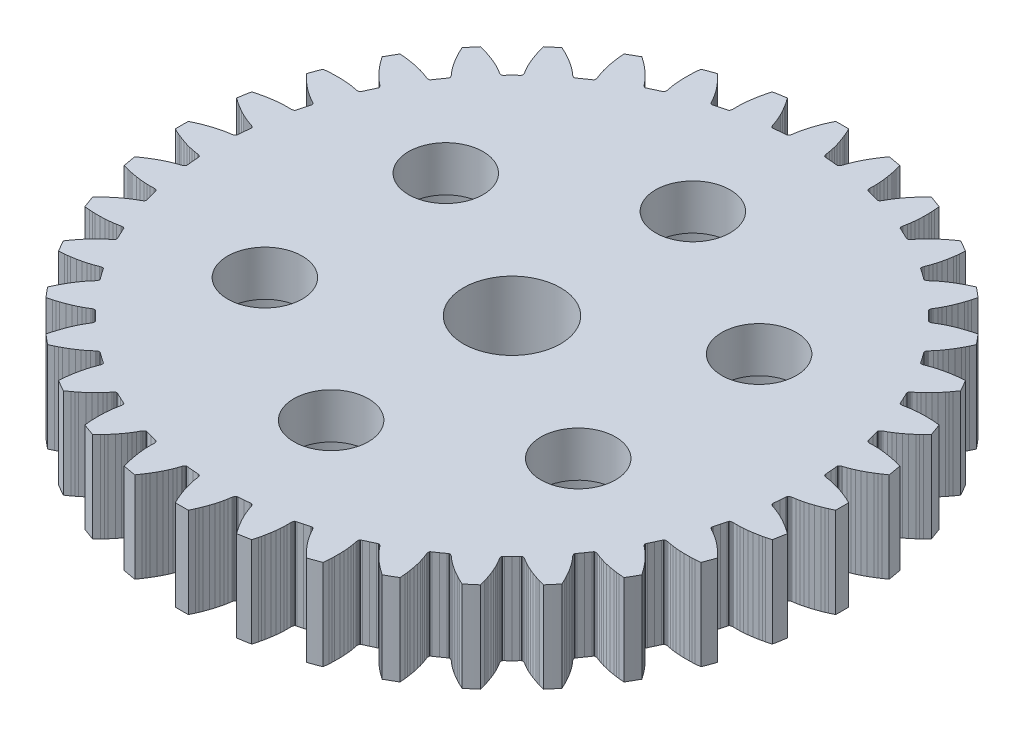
SolidWorks part; units mm, degrees
ref_plane "Front Plane" through (0, 0, 0) normal (0, 0, 1) x (1, 0, 0)
ref_plane "Top Plane" through (0, 0, 0) normal (0, 1, 0) x (1, 0, 0)
ref_plane "Right Plane" through (0, 0, 0) normal (1, 0, 0) x (0, 0, -1)
sketch "Sketch2" plane through (0, 0, 0) normal (0, 1, 0) x (1, 0, 0)
  line L632 (14.2382, 2.1155) -> (14.1321, 2.046)
  line L633 (14.1321, 2.046) -> (14.0302, 1.9822)
  line L634 (14.0302, 1.9822) -> (13.8362, 1.869)
  line L635 (13.8362, 1.869) -> (13.6574, 1.7744)
  line L636 (13.6574, 1.7744) -> (13.4969, 1.698)
  line L637 (13.4969, 1.698) -> (13.3538, 1.637)
  line L638 (13.3538, 1.637) -> (13.2277, 1.5894)
  line L639 (13.2277, 1.5894) -> (13.0788, 1.5394)
  line L640 (13.0788, 1.5394) -> (13.0417, 1.5232)
  line L641 (13.0417, 1.5232) -> (13.011, 1.5062)
  line L642 (13.011, 1.5062) -> (12.9867, 1.4887)
  line L643 (12.9867, 1.4887) -> (12.9688, 1.471)
  line L644 (12.9688, 1.471) -> (12.9574, 1.4533)
  line L645 (12.9574, 1.4533) -> (12.9524, 1.4359)
  line L646 (12.9524, 1.4359) -> (12.9583, 1.3725)
  line L647 (12.9583, 1.3725) -> (12.9811, 1.1357)
  line L648 (12.9811, 1.1357) -> (12.9998, 0.8985)
  line L649 (12.9998, 0.8985) -> (13.005, 0.8351)
  line L650 (13.005, 0.8351) -> (13.0129, 0.8188)
  line L651 (13.0129, 0.8188) -> (13.0272, 0.8034)
  line L652 (13.0272, 0.8034) -> (13.0479, 0.789)
  line L653 (13.0479, 0.789) -> (13.0749, 0.776)
  line L654 (13.0749, 0.776) -> (13.108, 0.7646)
  line L655 (13.108, 0.7646) -> (13.1474, 0.7551)
  line L656 (13.1474, 0.7551) -> (13.3028, 0.7317)
  line L657 (13.3028, 0.7317) -> (13.4352, 0.7067)
  line L658 (13.4352, 0.7067) -> (13.5867, 0.6715)
  line L659 (13.5867, 0.6715) -> (13.7581, 0.6241)
  line L660 (13.7581, 0.6241) -> (13.9505, 0.5621)
  line L662 (14.1613, 0.4843) -> (14.2727, 0.4391)
  line L663 (14.2727, 0.4391) -> (14.3893, 0.389)
  line L664 (14.3893, 0.389) -> (14.6039, 0.2893)
  line L665 (14.6039, -0.2893) -> (14.3893, -0.389)
  line L666 (14.3893, -0.389) -> (14.2727, -0.4391)
  line L667 (14.2727, -0.4391) -> (14.1613, -0.4843)
  line L668 (14.1613, -0.4843) -> (13.9505, -0.5621)
  line L669 (13.9505, -0.5621) -> (13.7581, -0.6241)
  line L670 (13.7581, -0.6241) -> (13.5867, -0.6715)
  line L671 (13.5867, -0.6715) -> (13.4352, -0.7067)
  line L672 (13.4352, -0.7067) -> (13.3028, -0.7317)
  line L673 (13.3028, -0.7317) -> (13.1474, -0.7551)
  line L674 (13.1474, -0.7551) -> (13.108, -0.7646)
  line L675 (13.108, -0.7646) -> (13.0749, -0.776)
  line L676 (13.0749, -0.776) -> (13.0479, -0.789)
  line L677 (13.0479, -0.789) -> (13.0272, -0.8034)
  line L678 (13.0272, -0.8034) -> (13.0129, -0.8188)
  line L679 (13.0129, -0.8188) -> (13.005, -0.8351)
  line L680 (13.005, -0.8351) -> (12.9998, -0.8985)
  line L681 (12.9998, -0.8985) -> (12.9811, -1.1357)
  line L682 (12.9811, -1.1357) -> (12.9583, -1.3725)
  line L683 (12.9583, -1.3725) -> (12.9524, -1.4359)
  line L684 (12.9524, -1.4359) -> (12.9574, -1.4533)
  line L685 (12.9574, -1.4533) -> (12.9688, -1.471)
  line L686 (12.9688, -1.471) -> (12.9867, -1.4887)
  line L687 (12.9867, -1.4887) -> (13.011, -1.5062)
  line L688 (13.011, -1.5062) -> (13.0417, -1.5232)
  line L689 (13.0417, -1.5232) -> (13.0788, -1.5394)
  line L690 (13.0788, -1.5394) -> (13.2277, -1.5894)
  line L691 (13.2277, -1.5894) -> (13.3538, -1.637)
  line L692 (13.3538, -1.637) -> (13.4969, -1.698)
  line L693 (13.4969, -1.698) -> (13.6574, -1.7744)
  line L694 (13.6574, -1.7744) -> (13.8362, -1.869)
  line L695 (13.8362, -1.869) -> (14.0302, -1.9822)
  line L696 (14.0302, -1.9822) -> (14.1321, -2.046)
  line L697 (14.1321, -2.046) -> (14.2382, -2.1155)
  line L698 (14.2382, -2.1155) -> (14.4322, -2.2511)
  line L699 (14.3318, -2.8208) -> (14.1031, -2.8818)
  line L700 (14.1031, -2.8818) -> (13.9796, -2.9109)
  line L701 (13.9796, -2.9109) -> (13.862, -2.936)
  line L702 (13.862, -2.936) -> (13.641, -2.976)
  line L703 (13.641, -2.976) -> (13.4407, -3.0037)
  line L704 (13.4407, -3.0037) -> (13.2637, -3.0206)
  line L705 (13.2637, -3.0206) -> (13.1084, -3.029)
  line L706 (13.1084, -3.029) -> (12.9736, -3.0306)
  line L707 (12.9736, -3.0306) -> (12.8166, -3.0266)
  line L708 (12.8166, -3.0266) -> (12.7761, -3.0292)
  line L709 (12.7761, -3.0292) -> (12.7415, -3.0347)
  line L710 (12.7415, -3.0347) -> (12.7127, -3.0428)
  line L711 (12.7127, -3.0428) -> (12.6898, -3.0534)
  line L712 (12.6898, -3.0534) -> (12.6731, -3.0661)
  line L713 (12.6731, -3.0661) -> (12.6624, -3.0807)
  line L714 (12.6624, -3.0807) -> (12.6462, -3.1422)
  line L715 (12.6462, -3.1422) -> (12.5867, -3.3726)
  line L716 (12.5867, -3.3726) -> (12.5231, -3.6019)
  line L717 (12.5231, -3.6019) -> (12.5063, -3.6632)
  line L718 (12.5063, -3.6632) -> (12.5082, -3.6812)
  line L719 (12.5082, -3.6812) -> (12.5164, -3.7006)
  line L720 (12.5164, -3.7006) -> (12.5309, -3.7212)
  line L721 (12.5309, -3.7212) -> (12.5518, -3.7426)
  line L722 (12.5518, -3.7426) -> (12.5791, -3.7647)
  line L723 (12.5791, -3.7647) -> (12.6128, -3.7872)
  line L724 (12.6128, -3.7872) -> (12.7508, -3.8623)
  line L725 (12.7508, -3.8623) -> (12.8667, -3.931)
  line L726 (12.8667, -3.931) -> (12.997, -4.0159)
  line L727 (12.997, -4.0159) -> (13.1418, -4.1191)
  line L728 (13.1418, -4.1191) -> (13.3015, -4.2432)
  line L729 (13.3015, -4.2432) -> (13.4729, -4.3884)
  line L730 (13.4729, -4.3884) -> (13.5621, -4.4689)
  line L731 (13.5621, -4.4689) -> (13.6545, -4.5558)
  line L732 (13.6545, -4.5558) -> (13.8221, -4.723)
  line L733 (13.6242, -5.2666) -> (13.3884, -5.287)
  line L734 (13.3884, -5.287) -> (13.2618, -5.2942)
  line L735 (13.2618, -5.2942) -> (13.1416, -5.2985)
  line L736 (13.1416, -5.2985) -> (12.917, -5.2995)
  line L737 (12.917, -5.2995) -> (12.7149, -5.292)
  line L738 (12.7149, -5.292) -> (12.5376, -5.2779)
  line L739 (12.5376, -5.2779) -> (12.3833, -5.2592)
  line L740 (12.3833, -5.2592) -> (12.2503, -5.2374)
  line L741 (12.2503, -5.2374) -> (12.0963, -5.2062)
  line L742 (12.0963, -5.2062) -> (12.056, -5.2017)
  line L743 (12.056, -5.2017) -> (12.0209, -5.2011)
  line L744 (12.0209, -5.2011) -> (11.9911, -5.2041)
  line L745 (11.9911, -5.2041) -> (11.9668, -5.2105)
  line L746 (11.9668, -5.2105) -> (11.9481, -5.2201)
  line L747 (11.9481, -5.2201) -> (11.9351, -5.2327)
  line L748 (11.9351, -5.2327) -> (11.9085, -5.2905)
  line L749 (11.9085, -5.2905) -> (11.8099, -5.507)
  line L750 (11.8099, -5.507) -> (11.7074, -5.7218)
  line L751 (11.7074, -5.7218) -> (11.6802, -5.7793)
  line L752 (11.6802, -5.7793) -> (11.679, -5.7973)
  line L753 (11.679, -5.7973) -> (11.6836, -5.8179)
  line L754 (11.6836, -5.8179) -> (11.6943, -5.8406)
  line L755 (11.6943, -5.8406) -> (11.7112, -5.8654)
  line L756 (11.7112, -5.8654) -> (11.7342, -5.8918)
  line L757 (11.7342, -5.8918) -> (11.7636, -5.9198)
  line L758 (11.7636, -5.9198) -> (11.8864, -6.0177)
  line L759 (11.8864, -6.0177) -> (11.9886, -6.1056)
  line L760 (11.9886, -6.1056) -> (12.1022, -6.2118)
  line L761 (12.1022, -6.2118) -> (12.2269, -6.3385)
  line L762 (12.2269, -6.3385) -> (12.3626, -6.4885)
  line L763 (12.3626, -6.4885) -> (12.5061, -6.6612)
  line L764 (12.5061, -6.6612) -> (12.5801, -6.7561)
  line L765 (12.5801, -6.7561) -> (12.656, -6.8577)
  line L766 (12.656, -6.8577) -> (12.7919, -7.0514)
  line L767 (12.5027, -7.5524) -> (12.2669, -7.5315)
  line L768 (12.2669, -7.5315) -> (12.141, -7.5166)
  line L769 (12.141, -7.5166) -> (12.0219, -7.5)
  line L770 (12.0219, -7.5) -> (11.8005, -7.462)
  line L771 (11.8005, -7.462) -> (11.6028, -7.4195)
  line L772 (11.6028, -7.4195) -> (11.4307, -7.3749)
  line L773 (11.4307, -7.3749) -> (11.2819, -7.3297)
  line L774 (11.2819, -7.3297) -> (11.1547, -7.2851)
  line L775 (11.1547, -7.2851) -> (11.0085, -7.2276)
  line L776 (11.0085, -7.2276) -> (10.9696, -7.2162)
  line L777 (10.9696, -7.2162) -> (10.9351, -7.2095)
  line L778 (10.9351, -7.2095) -> (10.9053, -7.2073)
  line L779 (10.9053, -7.2073) -> (10.8802, -7.2094)
  line L780 (10.8802, -7.2094) -> (10.8601, -7.2156)
  line L781 (10.8601, -7.2156) -> (10.8451, -7.2257)
  line L782 (10.8451, -7.2257) -> (10.8089, -7.278)
  line L783 (10.8089, -7.278) -> (10.6742, -7.4741)
  line L784 (10.6742, -7.4741) -> (10.5359, -7.6678)
  line L785 (10.5359, -7.6678) -> (10.4992, -7.7197)
  line L786 (10.4992, -7.7197) -> (10.4948, -7.7373)
  line L787 (10.4948, -7.7373) -> (10.4959, -7.7583)
  line L788 (10.4959, -7.7583) -> (10.5025, -7.7826)
  line L789 (10.5025, -7.7826) -> (10.5147, -7.8099)
  line L790 (10.5147, -7.8099) -> (10.5328, -7.84)
  line L791 (10.5328, -7.84) -> (10.5569, -7.8726)
  line L792 (10.5569, -7.8726) -> (10.6608, -7.9904)
  line L793 (10.6608, -7.9904) -> (10.7463, -8.0946)
  line L794 (10.7463, -8.0946) -> (10.8397, -8.2189)
  line L795 (10.8397, -8.2189) -> (10.9405, -8.3654)
  line L796 (10.9405, -8.3654) -> (11.048, -8.5367)
  line L797 (11.048, -8.5367) -> (11.1594, -8.7317)
  line L798 (11.1594, -8.7317) -> (11.2158, -8.8379)
  line L799 (11.2158, -8.8379) -> (11.2729, -8.9512)
  line L800 (11.2729, -8.9512) -> (11.3731, -9.1656)
  line L801 (11.0013, -9.6088) -> (10.7727, -9.5473)
  line L802 (10.7727, -9.5473) -> (10.6513, -9.5107)
  line L803 (10.6513, -9.5107) -> (10.5369, -9.4736)
  line L804 (10.5369, -9.4736) -> (10.3254, -9.3978)
  line L805 (10.3254, -9.3978) -> (10.1381, -9.3216)
  line L806 (10.1381, -9.3216) -> (9.9764, -9.2478)
  line L807 (9.9764, -9.2478) -> (9.8377, -9.1774)
  line L808 (9.8377, -9.1774) -> (9.7202, -9.1114)
  line L809 (9.7202, -9.1114) -> (9.5862, -9.0294)
  line L810 (9.5862, -9.0294) -> (9.5499, -9.0114)
  line L811 (9.5499, -9.0114) -> (9.5171, -8.9988)
  line L812 (9.5171, -8.9988) -> (9.4881, -8.9915)
  line L813 (9.4881, -8.9915) -> (9.463, -8.9892)
  line L814 (9.463, -8.9892) -> (9.4421, -8.9918)
  line L815 (9.4421, -8.9918) -> (9.4256, -8.9992)
  line L816 (9.4256, -8.9992) -> (9.3809, -9.0444)
  line L817 (9.3809, -9.0444) -> (9.2141, -9.2141)
  line L818 (9.2141, -9.2141) -> (9.0444, -9.3809)
  line L819 (9.0444, -9.3809) -> (8.9992, -9.4256)
  line L820 (8.9992, -9.4256) -> (8.9918, -9.4421)
  line L821 (8.9918, -9.4421) -> (8.9892, -9.463)
  line L822 (8.9892, -9.463) -> (8.9915, -9.4881)
  line L823 (8.9915, -9.4881) -> (8.9988, -9.5171)
  line L824 (8.9988, -9.5171) -> (9.0114, -9.5499)
  line L825 (9.0114, -9.5499) -> (9.0294, -9.5862)
  line L826 (9.0294, -9.5862) -> (9.1114, -9.7202)
  line L827 (9.1114, -9.7202) -> (9.1774, -9.8377)
  line L828 (9.1774, -9.8377) -> (9.2478, -9.9764)
  line L829 (9.2478, -9.9764) -> (9.3216, -10.1381)
  line L830 (9.3216, -10.1381) -> (9.3978, -10.3254)
  line L831 (9.3978, -10.3254) -> (9.4736, -10.5369)
  line L832 (9.4736, -10.5369) -> (9.5107, -10.6513)
  line L833 (9.5107, -10.6513) -> (9.5473, -10.7727)
  line L834 (9.5473, -10.7727) -> (9.6088, -11.0013)
  line L835 (9.1656, -11.3731) -> (8.9512, -11.2729)
  line L836 (8.9512, -11.2729) -> (8.8379, -11.2158)
  line L837 (8.8379, -11.2158) -> (8.7317, -11.1594)
  line L838 (8.7317, -11.1594) -> (8.5367, -11.048)
  line L839 (8.5367, -11.048) -> (8.3654, -10.9405)
  line L840 (8.3654, -10.9405) -> (8.2189, -10.8397)
  line L841 (8.2189, -10.8397) -> (8.0946, -10.7463)
  line L842 (8.0946, -10.7463) -> (7.9904, -10.6608)
  line L843 (7.9904, -10.6608) -> (7.8726, -10.5569)
  line L844 (7.8726, -10.5569) -> (7.84, -10.5328)
  line L845 (7.84, -10.5328) -> (7.8099, -10.5147)
  line L846 (7.8099, -10.5147) -> (7.7826, -10.5025)
  line L847 (7.7826, -10.5025) -> (7.7583, -10.4959)
  line L848 (7.7583, -10.4959) -> (7.7373, -10.4948)
  line L849 (7.7373, -10.4948) -> (7.7197, -10.4992)
  line L850 (7.7197, -10.4992) -> (7.6678, -10.5359)
  line L851 (7.6678, -10.5359) -> (7.4741, -10.6742)
  line L852 (7.4741, -10.6742) -> (7.278, -10.8089)
  line L853 (7.278, -10.8089) -> (7.2257, -10.8451)
  line L854 (7.2257, -10.8451) -> (7.2156, -10.8601)
  line L855 (7.2156, -10.8601) -> (7.2094, -10.8802)
  line L856 (7.2094, -10.8802) -> (7.2073, -10.9053)
  line L857 (7.2073, -10.9053) -> (7.2095, -10.9351)
  line L858 (7.2095, -10.9351) -> (7.2162, -10.9696)
  line L859 (7.2162, -10.9696) -> (7.2276, -11.0085)
  line L860 (7.2276, -11.0085) -> (7.2851, -11.1547)
  line L861 (7.2851, -11.1547) -> (7.3297, -11.2819)
  line L862 (7.3297, -11.2819) -> (7.3749, -11.4307)
  line L863 (7.3749, -11.4307) -> (7.4195, -11.6028)
  line L864 (7.4195, -11.6028) -> (7.462, -11.8005)
  line L865 (7.462, -11.8005) -> (7.5, -12.0219)
  line L866 (7.5, -12.0219) -> (7.5166, -12.141)
  line L867 (7.5166, -12.141) -> (7.5315, -12.2669)
  line L868 (7.5315, -12.2669) -> (7.5524, -12.5027)
  line L869 (7.0514, -12.7919) -> (6.8577, -12.656)
  line L870 (6.8577, -12.656) -> (6.7561, -12.5801)
  line L871 (6.7561, -12.5801) -> (6.6612, -12.5061)
  line L872 (6.6612, -12.5061) -> (6.4885, -12.3626)
  line L873 (6.4885, -12.3626) -> (6.3385, -12.2269)
  line L874 (6.3385, -12.2269) -> (6.2118, -12.1022)
  line L875 (6.2118, -12.1022) -> (6.1056, -11.9886)
  line L876 (6.1056, -11.9886) -> (6.0177, -11.8864)
  line L877 (6.0177, -11.8864) -> (5.9198, -11.7636)
  line L878 (5.9198, -11.7636) -> (5.8918, -11.7342)
  line L879 (5.8918, -11.7342) -> (5.8654, -11.7112)
  line L880 (5.8654, -11.7112) -> (5.8406, -11.6943)
  line L881 (5.8406, -11.6943) -> (5.8179, -11.6836)
  line L882 (5.8179, -11.6836) -> (5.7973, -11.679)
  line L883 (5.7973, -11.679) -> (5.7793, -11.6802)
  line L884 (5.7793, -11.6802) -> (5.7218, -11.7074)
  line L885 (5.7218, -11.7074) -> (5.507, -11.8099)
  line L886 (5.507, -11.8099) -> (5.2905, -11.9085)
  line L887 (5.2905, -11.9085) -> (5.2327, -11.9351)
  line L888 (5.2327, -11.9351) -> (5.2201, -11.9481)
  line L889 (5.2201, -11.9481) -> (5.2105, -11.9668)
  line L890 (5.2105, -11.9668) -> (5.2041, -11.9911)
  line L891 (5.2041, -11.9911) -> (5.2011, -12.0209)
  line L892 (5.2011, -12.0209) -> (5.2017, -12.056)
  line L893 (5.2017, -12.056) -> (5.2062, -12.0963)
  line L894 (5.2062, -12.0963) -> (5.2374, -12.2503)
  line L895 (5.2374, -12.2503) -> (5.2592, -12.3833)
  line L896 (5.2592, -12.3833) -> (5.2779, -12.5376)
  line L897 (5.2779, -12.5376) -> (5.292, -12.7149)
  line L898 (5.292, -12.7149) -> (5.2995, -12.917)
  line L899 (5.2995, -12.917) -> (5.2985, -13.1416)
  line L900 (5.2985, -13.1416) -> (5.2942, -13.2618)
  line L901 (5.2942, -13.2618) -> (5.287, -13.3884)
  line L902 (5.287, -13.3884) -> (5.2666, -13.6242)
  line L903 (4.723, -13.8221) -> (4.5558, -13.6545)
  line L904 (4.5558, -13.6545) -> (4.4689, -13.5621)
  line L905 (4.4689, -13.5621) -> (4.3884, -13.4729)
  line L906 (4.3884, -13.4729) -> (4.2432, -13.3015)
  line L907 (4.2432, -13.3015) -> (4.1191, -13.1418)
  line L908 (4.1191, -13.1418) -> (4.0159, -12.997)
  line L909 (4.0159, -12.997) -> (3.931, -12.8667)
  line L910 (3.931, -12.8667) -> (3.8623, -12.7508)
  line L911 (3.8623, -12.7508) -> (3.7872, -12.6128)
  line L912 (3.7872, -12.6128) -> (3.7647, -12.5791)
  line L913 (3.7647, -12.5791) -> (3.7426, -12.5518)
  line L914 (3.7426, -12.5518) -> (3.7212, -12.5309)
  line L915 (3.7212, -12.5309) -> (3.7006, -12.5164)
  line L916 (3.7006, -12.5164) -> (3.6812, -12.5082)
  line L917 (3.6812, -12.5082) -> (3.6632, -12.5063)
  line L918 (3.6632, -12.5063) -> (3.6019, -12.5231)
  line L919 (3.6019, -12.5231) -> (3.3726, -12.5867)
  line L920 (3.3726, -12.5867) -> (3.1422, -12.6462)
  line L921 (3.1422, -12.6462) -> (3.0807, -12.6624)
  line L922 (3.0807, -12.6624) -> (3.0661, -12.6731)
  line L923 (3.0661, -12.6731) -> (3.0534, -12.6898)
  line L924 (3.0534, -12.6898) -> (3.0428, -12.7127)
  line L925 (3.0428, -12.7127) -> (3.0347, -12.7415)
  line L926 (3.0347, -12.7415) -> (3.0292, -12.7761)
  line L927 (3.0292, -12.7761) -> (3.0266, -12.8166)
  line L928 (3.0266, -12.8166) -> (3.0306, -12.9736)
  line L929 (3.0306, -12.9736) -> (3.029, -13.1084)
  line L930 (3.029, -13.1084) -> (3.0206, -13.2637)
  line L931 (3.0206, -13.2637) -> (3.0037, -13.4407)
  line L932 (3.0037, -13.4407) -> (2.976, -13.641)
  line L933 (2.976, -13.641) -> (2.936, -13.862)
  line L934 (2.936, -13.862) -> (2.9109, -13.9796)
  line L935 (2.9109, -13.9796) -> (2.8818, -14.1031)
  line L936 (2.8818, -14.1031) -> (2.8208, -14.3318)
  line L937 (2.2511, -14.4322) -> (2.1155, -14.2382)
  line L938 (2.1155, -14.2382) -> (2.046, -14.1321)
  line L939 (2.046, -14.1321) -> (1.9822, -14.0302)
  line L940 (1.9822, -14.0302) -> (1.869, -13.8362)
  line L941 (1.869, -13.8362) -> (1.7744, -13.6574)
  line L942 (1.7744, -13.6574) -> (1.698, -13.4969)
  line L943 (1.698, -13.4969) -> (1.637, -13.3538)
  line L944 (1.637, -13.3538) -> (1.5894, -13.2277)
  line L945 (1.5894, -13.2277) -> (1.5394, -13.0788)
  line L946 (1.5394, -13.0788) -> (1.5232, -13.0417)
  line L947 (1.5232, -13.0417) -> (1.5062, -13.011)
  line L948 (1.5062, -13.011) -> (1.4887, -12.9867)
  line L949 (1.4887, -12.9867) -> (1.471, -12.9688)
  line L950 (1.471, -12.9688) -> (1.4533, -12.9574)
  line L951 (1.4533, -12.9574) -> (1.4359, -12.9524)
  line L952 (1.4359, -12.9524) -> (1.3725, -12.9583)
  line L953 (1.3725, -12.9583) -> (1.1357, -12.9811)
  line L954 (1.1357, -12.9811) -> (0.8985, -12.9998)
  line L955 (0.8985, -12.9998) -> (0.8351, -13.005)
  line L956 (0.8351, -13.005) -> (0.8188, -13.0129)
  line L957 (0.8188, -13.0129) -> (0.8034, -13.0272)
  line L958 (0.8034, -13.0272) -> (0.789, -13.0479)
  line L959 (0.789, -13.0479) -> (0.776, -13.0749)
  line L960 (0.776, -13.0749) -> (0.7646, -13.108)
  line L961 (0.7646, -13.108) -> (0.7551, -13.1474)
  line L962 (0.7551, -13.1474) -> (0.7317, -13.3028)
  line L963 (0.7317, -13.3028) -> (0.7067, -13.4352)
  line L964 (0.7067, -13.4352) -> (0.6715, -13.5867)
  line L965 (0.6715, -13.5867) -> (0.6241, -13.7581)
  line L966 (0.6241, -13.7581) -> (0.5621, -13.9505)
  line L967 (0.5621, -13.9505) -> (0.4843, -14.1613)
  line L968 (0.4843, -14.1613) -> (0.4391, -14.2727)
  line L969 (0.4391, -14.2727) -> (0.389, -14.3893)
  line L970 (0.389, -14.3893) -> (0.2893, -14.6039)
  line L971 (-0.2893, -14.6039) -> (-0.389, -14.3893)
  line L972 (-0.389, -14.3893) -> (-0.4391, -14.2727)
  line L973 (-0.4391, -14.2727) -> (-0.4843, -14.1613)
  line L974 (-0.4843, -14.1613) -> (-0.5621, -13.9505)
  line L975 (-0.5621, -13.9505) -> (-0.6241, -13.7581)
  line L976 (-0.6241, -13.7581) -> (-0.6715, -13.5867)
  line L977 (-0.6715, -13.5867) -> (-0.7067, -13.4352)
  line L978 (-0.7067, -13.4352) -> (-0.7317, -13.3028)
  line L979 (-0.7317, -13.3028) -> (-0.7551, -13.1474)
  line L980 (-0.7551, -13.1474) -> (-0.7646, -13.108)
  line L981 (-0.7646, -13.108) -> (-0.776, -13.0749)
  line L982 (-0.776, -13.0749) -> (-0.789, -13.0479)
  line L983 (-0.789, -13.0479) -> (-0.8034, -13.0272)
  line L984 (-0.8034, -13.0272) -> (-0.8188, -13.0129)
  line L985 (-0.8188, -13.0129) -> (-0.8351, -13.005)
  line L986 (-0.8351, -13.005) -> (-0.8985, -12.9998)
  line L987 (-0.8985, -12.9998) -> (-1.1357, -12.9811)
  line L988 (-1.1357, -12.9811) -> (-1.3725, -12.9583)
  line L989 (-1.3725, -12.9583) -> (-1.4359, -12.9524)
  line L990 (-1.4359, -12.9524) -> (-1.4533, -12.9574)
  line L991 (-1.4533, -12.9574) -> (-1.471, -12.9688)
  line L992 (-1.471, -12.9688) -> (-1.4887, -12.9867)
  line L993 (-1.4887, -12.9867) -> (-1.5062, -13.011)
  line L994 (-1.5062, -13.011) -> (-1.5232, -13.0417)
  line L995 (-1.5232, -13.0417) -> (-1.5394, -13.0788)
  line L996 (-1.5394, -13.0788) -> (-1.5894, -13.2277)
  line L997 (-1.5894, -13.2277) -> (-1.637, -13.3538)
  line L998 (-1.637, -13.3538) -> (-1.698, -13.4969)
  line L999 (-1.698, -13.4969) -> (-1.7744, -13.6574)
  line L1000 (-1.7744, -13.6574) -> (-1.869, -13.8362)
  line L1001 (-1.869, -13.8362) -> (-1.9822, -14.0302)
  line L1002 (-1.9822, -14.0302) -> (-2.046, -14.1321)
  line L1003 (-2.046, -14.1321) -> (-2.1155, -14.2382)
  line L1004 (-2.1155, -14.2382) -> (-2.2511, -14.4322)
  line L1005 (-2.8208, -14.3318) -> (-2.8818, -14.1031)
  line L1006 (-2.8818, -14.1031) -> (-2.9109, -13.9796)
  line L1007 (-2.9109, -13.9796) -> (-2.936, -13.862)
  line L1008 (-2.936, -13.862) -> (-2.976, -13.641)
  line L1009 (-2.976, -13.641) -> (-3.0037, -13.4407)
  line L1010 (-3.0037, -13.4407) -> (-3.0206, -13.2637)
  line L1011 (-3.0206, -13.2637) -> (-3.029, -13.1084)
  line L1012 (-3.029, -13.1084) -> (-3.0306, -12.9736)
  line L1013 (-3.0306, -12.9736) -> (-3.0266, -12.8166)
  line L1014 (-3.0266, -12.8166) -> (-3.0292, -12.7761)
  line L1015 (-3.0292, -12.7761) -> (-3.0347, -12.7415)
  line L1016 (-3.0347, -12.7415) -> (-3.0428, -12.7127)
  line L1017 (-3.0428, -12.7127) -> (-3.0534, -12.6898)
  line L1018 (-3.0534, -12.6898) -> (-3.0661, -12.6731)
  line L1019 (-3.0661, -12.6731) -> (-3.0807, -12.6624)
  line L1020 (-3.0807, -12.6624) -> (-3.1422, -12.6462)
  line L1021 (-3.1422, -12.6462) -> (-3.3726, -12.5867)
  line L1022 (-3.3726, -12.5867) -> (-3.6019, -12.5231)
  line L1023 (-3.6019, -12.5231) -> (-3.6632, -12.5063)
  line L1024 (-3.6632, -12.5063) -> (-3.6812, -12.5082)
  line L1025 (-3.6812, -12.5082) -> (-3.7006, -12.5164)
  line L1026 (-3.7006, -12.5164) -> (-3.7212, -12.5309)
  line L1027 (-3.7212, -12.5309) -> (-3.7426, -12.5518)
  line L1028 (-3.7426, -12.5518) -> (-3.7647, -12.5791)
  line L1029 (-3.7647, -12.5791) -> (-3.7872, -12.6128)
  line L1030 (-3.7872, -12.6128) -> (-3.8623, -12.7508)
  line L1031 (-3.8623, -12.7508) -> (-3.931, -12.8667)
  line L1032 (-3.931, -12.8667) -> (-4.0159, -12.997)
  line L1033 (-4.0159, -12.997) -> (-4.1191, -13.1418)
  line L1034 (-4.1191, -13.1418) -> (-4.2432, -13.3015)
  line L1035 (-4.2432, -13.3015) -> (-4.3884, -13.4729)
  line L1036 (-4.3884, -13.4729) -> (-4.4689, -13.5621)
  line L1037 (-4.4689, -13.5621) -> (-4.5558, -13.6545)
  line L1038 (-4.5558, -13.6545) -> (-4.723, -13.8221)
  line L1039 (-5.2666, -13.6242) -> (-5.287, -13.3884)
  line L1040 (-5.287, -13.3884) -> (-5.2942, -13.2618)
  line L1041 (-5.2942, -13.2618) -> (-5.2985, -13.1416)
  line L1042 (-5.2985, -13.1416) -> (-5.2995, -12.917)
  line L1043 (-5.2995, -12.917) -> (-5.292, -12.7149)
  line L1044 (-5.292, -12.7149) -> (-5.2779, -12.5376)
  line L1045 (-5.2779, -12.5376) -> (-5.2592, -12.3833)
  line L1046 (-5.2592, -12.3833) -> (-5.2374, -12.2503)
  line L1047 (-5.2374, -12.2503) -> (-5.2062, -12.0963)
  line L1048 (-5.2062, -12.0963) -> (-5.2017, -12.056)
  line L1049 (-5.2017, -12.056) -> (-5.2011, -12.0209)
  line L1050 (-5.2011, -12.0209) -> (-5.2041, -11.9911)
  line L1051 (-5.2041, -11.9911) -> (-5.2105, -11.9668)
  line L1052 (-5.2105, -11.9668) -> (-5.2201, -11.9481)
  line L1053 (-5.2201, -11.9481) -> (-5.2327, -11.9351)
  line L1054 (-5.2327, -11.9351) -> (-5.2905, -11.9085)
  line L1055 (-5.2905, -11.9085) -> (-5.507, -11.8099)
  line L1056 (-5.507, -11.8099) -> (-5.7218, -11.7074)
  line L1057 (-5.7218, -11.7074) -> (-5.7793, -11.6802)
  line L1058 (-5.7793, -11.6802) -> (-5.7973, -11.679)
  line L1059 (-5.7973, -11.679) -> (-5.8179, -11.6836)
  line L1060 (-5.8179, -11.6836) -> (-5.8406, -11.6943)
  line L1061 (-5.8406, -11.6943) -> (-5.8654, -11.7112)
  line L1062 (-5.8654, -11.7112) -> (-5.8918, -11.7342)
  line L1063 (-5.8918, -11.7342) -> (-5.9198, -11.7636)
  line L1064 (-5.9198, -11.7636) -> (-6.0177, -11.8864)
  line L1065 (-6.0177, -11.8864) -> (-6.1056, -11.9886)
  line L1066 (-6.1056, -11.9886) -> (-6.2118, -12.1022)
  line L1067 (-6.2118, -12.1022) -> (-6.3385, -12.2269)
  line L1068 (-6.3385, -12.2269) -> (-6.4885, -12.3626)
  line L1069 (-6.4885, -12.3626) -> (-6.6612, -12.5061)
  line L1070 (-6.6612, -12.5061) -> (-6.7561, -12.5801)
  line L1071 (-6.7561, -12.5801) -> (-6.8577, -12.656)
  line L1072 (-6.8577, -12.656) -> (-7.0514, -12.7919)
  line L1073 (-7.5524, -12.5027) -> (-7.5315, -12.2669)
  line L1074 (-7.5315, -12.2669) -> (-7.5166, -12.141)
  line L1075 (-7.5166, -12.141) -> (-7.5, -12.0219)
  line L1076 (-7.5, -12.0219) -> (-7.462, -11.8005)
  line L1077 (-7.462, -11.8005) -> (-7.4195, -11.6028)
  line L1078 (-7.4195, -11.6028) -> (-7.3749, -11.4307)
  line L1079 (-7.3749, -11.4307) -> (-7.3297, -11.2819)
  line L1080 (-7.3297, -11.2819) -> (-7.2851, -11.1547)
  line L1081 (-7.2851, -11.1547) -> (-7.2276, -11.0085)
  line L1082 (-7.2276, -11.0085) -> (-7.2162, -10.9696)
  line L1083 (-7.2162, -10.9696) -> (-7.2095, -10.9351)
  line L1084 (-7.2095, -10.9351) -> (-7.2073, -10.9053)
  line L1085 (-7.2073, -10.9053) -> (-7.2094, -10.8802)
  line L1086 (-7.2094, -10.8802) -> (-7.2156, -10.8601)
  line L1087 (-7.2156, -10.8601) -> (-7.2257, -10.8451)
  line L1088 (-7.2257, -10.8451) -> (-7.278, -10.8089)
  line L1089 (-7.278, -10.8089) -> (-7.4741, -10.6742)
  line L1090 (-7.4741, -10.6742) -> (-7.6678, -10.5359)
  line L1091 (-7.6678, -10.5359) -> (-7.7197, -10.4992)
  line L1092 (-7.7197, -10.4992) -> (-7.7373, -10.4948)
  line L1093 (-7.7373, -10.4948) -> (-7.7583, -10.4959)
  line L1094 (-7.7583, -10.4959) -> (-7.7826, -10.5025)
  line L1095 (-7.7826, -10.5025) -> (-7.8099, -10.5147)
  line L1096 (-7.8099, -10.5147) -> (-7.84, -10.5328)
  line L1097 (-7.84, -10.5328) -> (-7.8726, -10.5569)
  line L1098 (-7.8726, -10.5569) -> (-7.9904, -10.6608)
  line L1099 (-7.9904, -10.6608) -> (-8.0946, -10.7463)
  line L1100 (-8.0946, -10.7463) -> (-8.2189, -10.8397)
  line L1101 (-8.2189, -10.8397) -> (-8.3654, -10.9405)
  line L1102 (-8.3654, -10.9405) -> (-8.5367, -11.048)
  line L1103 (-8.5367, -11.048) -> (-8.7317, -11.1594)
  line L1104 (-8.7317, -11.1594) -> (-8.8379, -11.2158)
  line L1105 (-8.8379, -11.2158) -> (-8.9512, -11.2729)
  line L1106 (-8.9512, -11.2729) -> (-9.1656, -11.3731)
  line L1107 (-9.6088, -11.0013) -> (-9.5473, -10.7727)
  line L1108 (-9.5473, -10.7727) -> (-9.5107, -10.6513)
  line L1109 (-9.5107, -10.6513) -> (-9.4736, -10.5369)
  line L1110 (-9.4736, -10.5369) -> (-9.3978, -10.3254)
  line L1111 (-9.3978, -10.3254) -> (-9.3216, -10.1381)
  line L1112 (-9.3216, -10.1381) -> (-9.2478, -9.9764)
  line L1113 (-9.2478, -9.9764) -> (-9.1774, -9.8377)
  line L1114 (-9.1774, -9.8377) -> (-9.1114, -9.7202)
  line L1115 (-9.1114, -9.7202) -> (-9.0294, -9.5862)
  line L1116 (-9.0294, -9.5862) -> (-9.0114, -9.5499)
  line L1117 (-9.0114, -9.5499) -> (-8.9988, -9.5171)
  line L1118 (-8.9988, -9.5171) -> (-8.9915, -9.4881)
  line L1119 (-8.9915, -9.4881) -> (-8.9892, -9.463)
  line L1120 (-8.9892, -9.463) -> (-8.9918, -9.4421)
  line L1121 (-8.9918, -9.4421) -> (-8.9992, -9.4256)
  line L1122 (-8.9992, -9.4256) -> (-9.0444, -9.3809)
  line L1123 (-9.0444, -9.3809) -> (-9.2141, -9.2141)
  line L1124 (-9.2141, -9.2141) -> (-9.3809, -9.0444)
  line L1125 (-9.3809, -9.0444) -> (-9.4256, -8.9992)
  line L1126 (-9.4256, -8.9992) -> (-9.4421, -8.9918)
  line L1127 (-9.4421, -8.9918) -> (-9.463, -8.9892)
  line L1128 (-9.463, -8.9892) -> (-9.4881, -8.9915)
  line L1129 (-9.4881, -8.9915) -> (-9.5171, -8.9988)
  line L1130 (-9.5171, -8.9988) -> (-9.5499, -9.0114)
  line L1131 (-9.5499, -9.0114) -> (-9.5862, -9.0294)
  line L1132 (-9.5862, -9.0294) -> (-9.7202, -9.1114)
  line L1133 (-9.7202, -9.1114) -> (-9.8377, -9.1774)
  line L1134 (-9.8377, -9.1774) -> (-9.9764, -9.2478)
  line L1135 (-9.9764, -9.2478) -> (-10.1381, -9.3216)
  line L1136 (-10.1381, -9.3216) -> (-10.3254, -9.3978)
  line L1137 (-10.3254, -9.3978) -> (-10.5369, -9.4736)
  line L1138 (-10.5369, -9.4736) -> (-10.6513, -9.5107)
  line L1139 (-10.6513, -9.5107) -> (-10.7727, -9.5473)
  line L1140 (-10.7727, -9.5473) -> (-11.0013, -9.6088)
  line L1141 (-11.3731, -9.1656) -> (-11.2729, -8.9512)
  line L1142 (-11.2729, -8.9512) -> (-11.2158, -8.8379)
  line L1143 (-11.2158, -8.8379) -> (-11.1594, -8.7317)
  line L1144 (-11.1594, -8.7317) -> (-11.048, -8.5367)
  line L1145 (-11.048, -8.5367) -> (-10.9405, -8.3654)
  line L1146 (-10.9405, -8.3654) -> (-10.8397, -8.2189)
  line L1147 (-10.8397, -8.2189) -> (-10.7463, -8.0946)
  line L1148 (-10.7463, -8.0946) -> (-10.6608, -7.9904)
  line L1149 (-10.6608, -7.9904) -> (-10.5569, -7.8726)
  line L1150 (-10.5569, -7.8726) -> (-10.5328, -7.84)
  line L1151 (-10.5328, -7.84) -> (-10.5147, -7.8099)
  line L1152 (-10.5147, -7.8099) -> (-10.5025, -7.7826)
  line L1153 (-10.5025, -7.7826) -> (-10.4959, -7.7583)
  line L1154 (-10.4959, -7.7583) -> (-10.4948, -7.7373)
  line L1155 (-10.4948, -7.7373) -> (-10.4992, -7.7197)
  line L1156 (-10.4992, -7.7197) -> (-10.5359, -7.6678)
  line L1157 (-10.5359, -7.6678) -> (-10.6742, -7.4741)
  line L1158 (-10.6742, -7.4741) -> (-10.8089, -7.278)
  line L1159 (-10.8089, -7.278) -> (-10.8451, -7.2257)
  line L1160 (-10.8451, -7.2257) -> (-10.8601, -7.2156)
  line L1161 (-10.8601, -7.2156) -> (-10.8802, -7.2094)
  line L1162 (-10.8802, -7.2094) -> (-10.9053, -7.2073)
  line L1163 (-10.9053, -7.2073) -> (-10.9351, -7.2095)
  line L1164 (-10.9351, -7.2095) -> (-10.9696, -7.2162)
  line L1165 (-10.9696, -7.2162) -> (-11.0085, -7.2276)
  line L1166 (-11.0085, -7.2276) -> (-11.1547, -7.2851)
  line L1167 (-11.1547, -7.2851) -> (-11.2819, -7.3297)
  line L1168 (-11.2819, -7.3297) -> (-11.4307, -7.3749)
  line L1169 (-11.4307, -7.3749) -> (-11.6028, -7.4195)
  line L1170 (-11.6028, -7.4195) -> (-11.8005, -7.462)
  line L1171 (-11.8005, -7.462) -> (-12.0219, -7.5)
  line L1172 (-12.0219, -7.5) -> (-12.141, -7.5166)
  line L1173 (-12.141, -7.5166) -> (-12.2669, -7.5315)
  line L1174 (-12.2669, -7.5315) -> (-12.5027, -7.5524)
  line L1175 (-12.7919, -7.0514) -> (-12.656, -6.8577)
  line L1176 (-12.656, -6.8577) -> (-12.5801, -6.7561)
  line L1177 (-12.5801, -6.7561) -> (-12.5061, -6.6612)
  line L1178 (-12.5061, -6.6612) -> (-12.3626, -6.4885)
  line L1179 (-12.3626, -6.4885) -> (-12.2269, -6.3385)
  line L1180 (-12.2269, -6.3385) -> (-12.1022, -6.2118)
  line L1181 (-12.1022, -6.2118) -> (-11.9886, -6.1056)
  line L1182 (-11.9886, -6.1056) -> (-11.8864, -6.0177)
  line L1183 (-11.8864, -6.0177) -> (-11.7636, -5.9198)
  line L1184 (-11.7636, -5.9198) -> (-11.7342, -5.8918)
  line L1185 (-11.7342, -5.8918) -> (-11.7112, -5.8654)
  line L1186 (-11.7112, -5.8654) -> (-11.6943, -5.8406)
  line L1187 (-11.6943, -5.8406) -> (-11.6836, -5.8179)
  line L1188 (-11.6836, -5.8179) -> (-11.679, -5.7973)
  line L1189 (-11.679, -5.7973) -> (-11.6802, -5.7793)
  line L1190 (-11.6802, -5.7793) -> (-11.7074, -5.7218)
  line L1191 (-11.7074, -5.7218) -> (-11.8099, -5.507)
  line L1192 (-11.8099, -5.507) -> (-11.9085, -5.2905)
  line L1193 (-11.9085, -5.2905) -> (-11.9351, -5.2327)
  line L1194 (-11.9351, -5.2327) -> (-11.9481, -5.2201)
  line L1195 (-11.9481, -5.2201) -> (-11.9668, -5.2105)
  line L1196 (-11.9668, -5.2105) -> (-11.9911, -5.2041)
  line L1197 (-11.9911, -5.2041) -> (-12.0209, -5.2011)
  line L1198 (-12.0209, -5.2011) -> (-12.056, -5.2017)
  line L1199 (-12.056, -5.2017) -> (-12.0963, -5.2062)
  line L1200 (-12.0963, -5.2062) -> (-12.2503, -5.2374)
  line L1201 (-12.2503, -5.2374) -> (-12.3833, -5.2592)
  line L1202 (-12.3833, -5.2592) -> (-12.5376, -5.2779)
  line L1203 (-12.5376, -5.2779) -> (-12.7149, -5.292)
  line L1204 (-12.7149, -5.292) -> (-12.917, -5.2995)
  line L1205 (-12.917, -5.2995) -> (-13.1416, -5.2985)
  line L1206 (-13.1416, -5.2985) -> (-13.2618, -5.2942)
  line L1207 (-13.2618, -5.2942) -> (-13.3884, -5.287)
  line L1208 (-13.3884, -5.287) -> (-13.6242, -5.2666)
  line L1209 (-13.8221, -4.723) -> (-13.6545, -4.5558)
  line L1210 (-13.6545, -4.5558) -> (-13.5621, -4.4689)
  line L1211 (-13.5621, -4.4689) -> (-13.4729, -4.3884)
  line L1212 (-13.4729, -4.3884) -> (-13.3015, -4.2432)
  line L1213 (-13.3015, -4.2432) -> (-13.1418, -4.1191)
  line L1214 (-13.1418, -4.1191) -> (-12.997, -4.0159)
  line L1215 (-12.997, -4.0159) -> (-12.8667, -3.931)
  line L1216 (-12.8667, -3.931) -> (-12.7508, -3.8623)
  line L1217 (-12.7508, -3.8623) -> (-12.6128, -3.7872)
  line L1218 (-12.6128, -3.7872) -> (-12.5791, -3.7647)
  line L1219 (-12.5791, -3.7647) -> (-12.5518, -3.7426)
  line L1220 (-12.5518, -3.7426) -> (-12.5309, -3.7212)
  line L1221 (-12.5309, -3.7212) -> (-12.5164, -3.7006)
  line L1222 (-12.5164, -3.7006) -> (-12.5082, -3.6812)
  line L1223 (-12.5082, -3.6812) -> (-12.5063, -3.6632)
  line L1224 (-12.5063, -3.6632) -> (-12.5231, -3.6019)
  line L1225 (-12.5231, -3.6019) -> (-12.5867, -3.3726)
  line L1226 (-12.5867, -3.3726) -> (-12.6462, -3.1422)
  line L1227 (-12.6462, -3.1422) -> (-12.6624, -3.0807)
  line L1228 (-12.6624, -3.0807) -> (-12.6731, -3.0661)
  line L1229 (-12.6731, -3.0661) -> (-12.6898, -3.0534)
  line L1230 (-12.6898, -3.0534) -> (-12.7127, -3.0428)
  line L1231 (-12.7127, -3.0428) -> (-12.7415, -3.0347)
  line L1232 (-12.7415, -3.0347) -> (-12.7761, -3.0292)
  line L1233 (-12.7761, -3.0292) -> (-12.8166, -3.0266)
  line L1234 (-12.8166, -3.0266) -> (-12.9736, -3.0306)
  line L1235 (-12.9736, -3.0306) -> (-13.1084, -3.029)
  line L1236 (-13.1084, -3.029) -> (-13.2637, -3.0206)
  line L1237 (-13.2637, -3.0206) -> (-13.4407, -3.0037)
  line L1238 (-13.4407, -3.0037) -> (-13.641, -2.976)
  line L1239 (-13.641, -2.976) -> (-13.862, -2.936)
  line L1240 (-13.862, -2.936) -> (-13.9796, -2.9109)
  line L1241 (-13.9796, -2.9109) -> (-14.1031, -2.8818)
  line L1242 (-14.1031, -2.8818) -> (-14.3318, -2.8208)
  line L1243 (-14.4322, -2.2511) -> (-14.2382, -2.1155)
  line L1244 (-14.2382, -2.1155) -> (-14.1321, -2.046)
  line L1245 (-14.1321, -2.046) -> (-14.0302, -1.9822)
  line L1246 (-14.0302, -1.9822) -> (-13.8362, -1.869)
  line L1247 (-13.8362, -1.869) -> (-13.6574, -1.7744)
  line L1248 (-13.6574, -1.7744) -> (-13.4969, -1.698)
  line L1249 (-13.4969, -1.698) -> (-13.3538, -1.637)
  line L1250 (-13.3538, -1.637) -> (-13.2277, -1.5894)
  line L1251 (-13.2277, -1.5894) -> (-13.0788, -1.5394)
  line L1252 (-13.0788, -1.5394) -> (-13.0417, -1.5232)
  line L1253 (-13.0417, -1.5232) -> (-13.011, -1.5062)
  line L1254 (-13.011, -1.5062) -> (-12.9867, -1.4887)
  line L1255 (-12.9867, -1.4887) -> (-12.9688, -1.471)
  line L1256 (-12.9688, -1.471) -> (-12.9574, -1.4533)
  line L1257 (-12.9574, -1.4533) -> (-12.9524, -1.4359)
  line L1258 (-12.9524, -1.4359) -> (-12.9583, -1.3725)
  line L1259 (-12.9583, -1.3725) -> (-12.9811, -1.1357)
  line L1260 (-12.9811, -1.1357) -> (-12.9998, -0.8985)
  line L1261 (-12.9998, -0.8985) -> (-13.005, -0.8351)
  line L1262 (-13.005, -0.8351) -> (-13.0129, -0.8188)
  line L1263 (-13.0129, -0.8188) -> (-13.0272, -0.8034)
  line L1264 (-13.0272, -0.8034) -> (-13.0479, -0.789)
  line L1265 (-13.0479, -0.789) -> (-13.0749, -0.776)
  line L1266 (-13.0749, -0.776) -> (-13.108, -0.7646)
  line L1267 (-13.108, -0.7646) -> (-13.1474, -0.7551)
  line L1268 (-13.1474, -0.7551) -> (-13.3028, -0.7317)
  line L1269 (-13.3028, -0.7317) -> (-13.4352, -0.7067)
  line L1270 (-13.4352, -0.7067) -> (-13.5867, -0.6715)
  line L1271 (-13.5867, -0.6715) -> (-13.7581, -0.6241)
  line L1272 (-13.7581, -0.6241) -> (-13.9505, -0.5621)
  line L1273 (-13.9505, -0.5621) -> (-14.1613, -0.4843)
  line L1274 (-14.1613, -0.4843) -> (-14.2727, -0.4391)
  line L1275 (-14.2727, -0.4391) -> (-14.3893, -0.389)
  line L1276 (-14.3893, -0.389) -> (-14.6039, -0.2893)
  line L1277 (-14.6039, 0.2893) -> (-14.3893, 0.389)
  line L1278 (-14.3893, 0.389) -> (-14.2727, 0.4391)
  line L1279 (-14.2727, 0.4391) -> (-14.1613, 0.4843)
  line L1280 (-14.1613, 0.4843) -> (-13.9505, 0.5621)
  line L1281 (-13.9505, 0.5621) -> (-13.7581, 0.6241)
  line L1282 (-13.7581, 0.6241) -> (-13.5867, 0.6715)
  line L1283 (-13.5867, 0.6715) -> (-13.4352, 0.7067)
  line L1284 (-13.4352, 0.7067) -> (-13.3028, 0.7317)
  line L1285 (-13.3028, 0.7317) -> (-13.1474, 0.7551)
  line L1286 (-13.1474, 0.7551) -> (-13.108, 0.7646)
  line L1287 (-13.108, 0.7646) -> (-13.0749, 0.776)
  line L1288 (-13.0749, 0.776) -> (-13.0479, 0.789)
  line L1289 (-13.0479, 0.789) -> (-13.0272, 0.8034)
  line L1290 (-13.0272, 0.8034) -> (-13.0129, 0.8188)
  line L1291 (-13.0129, 0.8188) -> (-13.005, 0.8351)
  line L1292 (-13.005, 0.8351) -> (-12.9998, 0.8985)
  line L1293 (-12.9998, 0.8985) -> (-12.9811, 1.1357)
  line L1294 (-12.9811, 1.1357) -> (-12.9583, 1.3725)
  line L1295 (-12.9583, 1.3725) -> (-12.9524, 1.4359)
  line L1296 (-12.9524, 1.4359) -> (-12.9574, 1.4533)
  line L1297 (-12.9574, 1.4533) -> (-12.9688, 1.471)
  line L1298 (-12.9688, 1.471) -> (-12.9867, 1.4887)
  line L1299 (-12.9867, 1.4887) -> (-13.011, 1.5062)
  line L1300 (-13.011, 1.5062) -> (-13.0417, 1.5232)
  line L1301 (-13.0417, 1.5232) -> (-13.0788, 1.5394)
  line L1302 (-13.0788, 1.5394) -> (-13.2277, 1.5894)
  line L1303 (-13.2277, 1.5894) -> (-13.3538, 1.637)
  line L1304 (-13.3538, 1.637) -> (-13.4969, 1.698)
  line L1305 (-13.4969, 1.698) -> (-13.6574, 1.7744)
  line L1306 (-13.6574, 1.7744) -> (-13.8362, 1.869)
  line L1307 (-13.8362, 1.869) -> (-14.0302, 1.9822)
  line L1308 (-14.0302, 1.9822) -> (-14.1321, 2.046)
  line L1309 (-14.1321, 2.046) -> (-14.2382, 2.1155)
  line L1310 (-14.2382, 2.1155) -> (-14.4322, 2.2511)
  line L1311 (-14.3318, 2.8208) -> (-14.1031, 2.8818)
  line L1312 (-14.1031, 2.8818) -> (-13.9796, 2.9109)
  line L1313 (-13.9796, 2.9109) -> (-13.862, 2.936)
  line L1314 (-13.862, 2.936) -> (-13.641, 2.976)
  line L1315 (-13.641, 2.976) -> (-13.4407, 3.0037)
  line L1316 (-13.4407, 3.0037) -> (-13.2637, 3.0206)
  line L1317 (-13.2637, 3.0206) -> (-13.1084, 3.029)
  line L1318 (-13.1084, 3.029) -> (-12.9736, 3.0306)
  line L1319 (-12.9736, 3.0306) -> (-12.8166, 3.0266)
  line L1320 (-12.8166, 3.0266) -> (-12.7761, 3.0292)
  line L1321 (-12.7761, 3.0292) -> (-12.7415, 3.0347)
  line L1322 (-12.7415, 3.0347) -> (-12.7127, 3.0428)
  line L1323 (-12.7127, 3.0428) -> (-12.6898, 3.0534)
  line L1324 (-12.6898, 3.0534) -> (-12.6731, 3.0661)
  line L1325 (-12.6731, 3.0661) -> (-12.6624, 3.0807)
  line L1326 (-12.6624, 3.0807) -> (-12.6462, 3.1422)
  line L1327 (-12.6462, 3.1422) -> (-12.5867, 3.3726)
  line L1328 (-12.5867, 3.3726) -> (-12.5231, 3.6019)
  line L1329 (-12.5231, 3.6019) -> (-12.5063, 3.6632)
  line L1330 (-12.5063, 3.6632) -> (-12.5082, 3.6812)
  line L1331 (-12.5082, 3.6812) -> (-12.5164, 3.7006)
  line L1332 (-12.5164, 3.7006) -> (-12.5309, 3.7212)
  line L1333 (-12.5309, 3.7212) -> (-12.5518, 3.7426)
  line L1334 (-12.5518, 3.7426) -> (-12.5791, 3.7647)
  line L1335 (-12.5791, 3.7647) -> (-12.6128, 3.7872)
  line L1336 (-12.6128, 3.7872) -> (-12.7508, 3.8623)
  line L1337 (-12.7508, 3.8623) -> (-12.8667, 3.931)
  line L1338 (-12.8667, 3.931) -> (-12.997, 4.0159)
  line L1339 (-12.997, 4.0159) -> (-13.1418, 4.1191)
  line L1340 (-13.1418, 4.1191) -> (-13.3015, 4.2432)
  line L1341 (-13.3015, 4.2432) -> (-13.4729, 4.3884)
  line L1342 (-13.4729, 4.3884) -> (-13.5621, 4.4689)
  line L1343 (-13.5621, 4.4689) -> (-13.6545, 4.5558)
  line L1344 (-13.6545, 4.5558) -> (-13.8221, 4.723)
  line L1345 (-13.6242, 5.2666) -> (-13.3884, 5.287)
  line L1346 (-13.3884, 5.287) -> (-13.2618, 5.2942)
  line L1347 (-13.2618, 5.2942) -> (-13.1416, 5.2985)
  line L1348 (-13.1416, 5.2985) -> (-12.917, 5.2995)
  line L1349 (-12.917, 5.2995) -> (-12.7149, 5.292)
  line L1350 (-12.7149, 5.292) -> (-12.5376, 5.2779)
  line L1351 (-12.5376, 5.2779) -> (-12.3833, 5.2592)
  line L1352 (-12.3833, 5.2592) -> (-12.2503, 5.2374)
  line L1353 (-12.2503, 5.2374) -> (-12.0963, 5.2062)
  line L1354 (-12.0963, 5.2062) -> (-12.056, 5.2017)
  line L1355 (-12.056, 5.2017) -> (-12.0209, 5.2011)
  line L1356 (-12.0209, 5.2011) -> (-11.9911, 5.2041)
  line L1357 (-11.9911, 5.2041) -> (-11.9668, 5.2105)
  line L1358 (-11.9668, 5.2105) -> (-11.9481, 5.2201)
  line L1359 (-11.9481, 5.2201) -> (-11.9351, 5.2327)
  line L1360 (-11.9351, 5.2327) -> (-11.9085, 5.2905)
  line L1361 (-11.9085, 5.2905) -> (-11.8099, 5.507)
  line L1362 (-11.8099, 5.507) -> (-11.7074, 5.7218)
  line L1363 (-11.7074, 5.7218) -> (-11.6802, 5.7793)
  line L1364 (-11.6802, 5.7793) -> (-11.679, 5.7973)
  line L1365 (-11.679, 5.7973) -> (-11.6836, 5.8179)
  line L1366 (-11.6836, 5.8179) -> (-11.6943, 5.8406)
  line L1367 (-11.6943, 5.8406) -> (-11.7112, 5.8654)
  line L1368 (-11.7112, 5.8654) -> (-11.7342, 5.8918)
  line L1369 (-11.7342, 5.8918) -> (-11.7636, 5.9198)
  line L1370 (-11.7636, 5.9198) -> (-11.8864, 6.0177)
  line L1371 (-11.8864, 6.0177) -> (-11.9886, 6.1056)
  line L1372 (-11.9886, 6.1056) -> (-12.1022, 6.2118)
  line L1373 (-12.1022, 6.2118) -> (-12.2269, 6.3385)
  line L1374 (-12.2269, 6.3385) -> (-12.3626, 6.4885)
  line L1375 (-12.3626, 6.4885) -> (-12.5061, 6.6612)
  line L1376 (-12.5061, 6.6612) -> (-12.5801, 6.7561)
  line L1377 (-12.5801, 6.7561) -> (-12.656, 6.8577)
  line L1378 (-12.656, 6.8577) -> (-12.7919, 7.0514)
  line L1379 (-12.5027, 7.5524) -> (-12.2669, 7.5315)
  line L1380 (-12.2669, 7.5315) -> (-12.141, 7.5166)
  line L1381 (-12.141, 7.5166) -> (-12.0219, 7.5)
  line L1382 (-12.0219, 7.5) -> (-11.8005, 7.462)
  line L1383 (-11.8005, 7.462) -> (-11.6028, 7.4195)
  line L1384 (-11.6028, 7.4195) -> (-11.4307, 7.3749)
  line L1385 (-11.4307, 7.3749) -> (-11.2819, 7.3297)
  line L1386 (-11.2819, 7.3297) -> (-11.1547, 7.2851)
  line L1387 (-11.1547, 7.2851) -> (-11.0085, 7.2276)
  line L1388 (-11.0085, 7.2276) -> (-10.9696, 7.2162)
  line L1389 (-10.9696, 7.2162) -> (-10.9351, 7.2095)
  line L1390 (-10.9351, 7.2095) -> (-10.9053, 7.2073)
  line L1391 (-10.9053, 7.2073) -> (-10.8802, 7.2094)
  line L1392 (-10.8802, 7.2094) -> (-10.8601, 7.2156)
  line L1393 (-10.8601, 7.2156) -> (-10.8451, 7.2257)
  line L1394 (-10.8451, 7.2257) -> (-10.8089, 7.278)
  line L1395 (-10.8089, 7.278) -> (-10.6742, 7.4741)
  line L1396 (-10.6742, 7.4741) -> (-10.5359, 7.6678)
  line L1397 (-10.5359, 7.6678) -> (-10.4992, 7.7197)
  line L1398 (-10.4992, 7.7197) -> (-10.4948, 7.7373)
  line L1399 (-10.4948, 7.7373) -> (-10.4959, 7.7583)
  line L1400 (-10.4959, 7.7583) -> (-10.5025, 7.7826)
  line L1401 (-10.5025, 7.7826) -> (-10.5147, 7.8099)
  line L1402 (-10.5147, 7.8099) -> (-10.5328, 7.84)
  line L1403 (-10.5328, 7.84) -> (-10.5569, 7.8726)
  line L1404 (-10.5569, 7.8726) -> (-10.6608, 7.9904)
  line L1405 (-10.6608, 7.9904) -> (-10.7463, 8.0946)
  line L1406 (-10.7463, 8.0946) -> (-10.8397, 8.2189)
  line L1407 (-10.8397, 8.2189) -> (-10.9405, 8.3654)
  line L1408 (-10.9405, 8.3654) -> (-11.048, 8.5367)
  line L1409 (-11.048, 8.5367) -> (-11.1594, 8.7317)
  line L1410 (-11.1594, 8.7317) -> (-11.2158, 8.8379)
  line L1411 (-11.2158, 8.8379) -> (-11.2729, 8.9512)
  line L1412 (-11.2729, 8.9512) -> (-11.3731, 9.1656)
  line L1413 (-11.0013, 9.6088) -> (-10.7727, 9.5473)
  line L1414 (-10.7727, 9.5473) -> (-10.6513, 9.5107)
  line L1415 (-10.6513, 9.5107) -> (-10.5369, 9.4736)
  line L1416 (-10.5369, 9.4736) -> (-10.3254, 9.3978)
  line L1417 (-10.3254, 9.3978) -> (-10.1381, 9.3216)
  line L1418 (-10.1381, 9.3216) -> (-9.9764, 9.2478)
  line L1419 (-9.9764, 9.2478) -> (-9.8377, 9.1774)
  line L1420 (-9.8377, 9.1774) -> (-9.7202, 9.1114)
  line L1421 (-9.7202, 9.1114) -> (-9.5862, 9.0294)
  line L1422 (-9.5862, 9.0294) -> (-9.5499, 9.0114)
  line L1423 (-9.5499, 9.0114) -> (-9.5171, 8.9988)
  line L1424 (-9.5171, 8.9988) -> (-9.4881, 8.9915)
  line L1425 (-9.4881, 8.9915) -> (-9.463, 8.9892)
  line L1426 (-9.463, 8.9892) -> (-9.4421, 8.9918)
  line L1427 (-9.4421, 8.9918) -> (-9.4256, 8.9992)
  line L1428 (-9.4256, 8.9992) -> (-9.3809, 9.0444)
  line L1429 (-9.3809, 9.0444) -> (-9.2141, 9.2141)
  line L1430 (-9.2141, 9.2141) -> (-9.0444, 9.3809)
  line L1431 (-9.0444, 9.3809) -> (-8.9992, 9.4256)
  line L1432 (-8.9992, 9.4256) -> (-8.9918, 9.4421)
  line L1433 (-8.9918, 9.4421) -> (-8.9892, 9.463)
  line L1434 (-8.9892, 9.463) -> (-8.9915, 9.4881)
  line L1435 (-8.9915, 9.4881) -> (-8.9988, 9.5171)
  line L1436 (-8.9988, 9.5171) -> (-9.0114, 9.5499)
  line L1437 (-9.0114, 9.5499) -> (-9.0294, 9.5862)
  line L1438 (-9.0294, 9.5862) -> (-9.1114, 9.7202)
  line L1439 (-9.1114, 9.7202) -> (-9.1774, 9.8377)
  line L1440 (-9.1774, 9.8377) -> (-9.2478, 9.9764)
  line L1441 (-9.2478, 9.9764) -> (-9.3216, 10.1381)
  line L1442 (-9.3216, 10.1381) -> (-9.3978, 10.3254)
  line L1443 (-9.3978, 10.3254) -> (-9.4736, 10.5369)
  line L1444 (-9.4736, 10.5369) -> (-9.5107, 10.6513)
  line L1445 (-9.5107, 10.6513) -> (-9.5473, 10.7727)
  line L1446 (-9.5473, 10.7727) -> (-9.6088, 11.0013)
  line L1447 (-9.1656, 11.3731) -> (-8.9512, 11.2729)
  line L1448 (-8.9512, 11.2729) -> (-8.8379, 11.2158)
  line L1449 (-8.8379, 11.2158) -> (-8.7317, 11.1594)
  line L1450 (-8.7317, 11.1594) -> (-8.5367, 11.048)
  line L1451 (-8.5367, 11.048) -> (-8.3654, 10.9405)
  line L1452 (-8.3654, 10.9405) -> (-8.2189, 10.8397)
  line L1453 (-8.2189, 10.8397) -> (-8.0946, 10.7463)
  line L1454 (-8.0946, 10.7463) -> (-7.9904, 10.6608)
  line L1455 (-7.9904, 10.6608) -> (-7.8726, 10.5569)
  line L1456 (-7.8726, 10.5569) -> (-7.84, 10.5328)
  line L1457 (-7.84, 10.5328) -> (-7.8099, 10.5147)
  line L1458 (-7.8099, 10.5147) -> (-7.7826, 10.5025)
  line L1459 (-7.7826, 10.5025) -> (-7.7583, 10.4959)
  line L1460 (-7.7583, 10.4959) -> (-7.7373, 10.4948)
  line L1461 (-7.7373, 10.4948) -> (-7.7197, 10.4992)
  line L1462 (-7.7197, 10.4992) -> (-7.6678, 10.5359)
  line L1463 (-7.6678, 10.5359) -> (-7.4741, 10.6742)
  line L1464 (-7.4741, 10.6742) -> (-7.278, 10.8089)
  line L1465 (-7.278, 10.8089) -> (-7.2257, 10.8451)
  line L1466 (-7.2257, 10.8451) -> (-7.2156, 10.8601)
  line L1467 (-7.2156, 10.8601) -> (-7.2094, 10.8802)
  line L1468 (-7.2094, 10.8802) -> (-7.2073, 10.9053)
  line L1469 (-7.2073, 10.9053) -> (-7.2095, 10.9351)
  line L1470 (-7.2095, 10.9351) -> (-7.2162, 10.9696)
  line L1471 (-7.2162, 10.9696) -> (-7.2276, 11.0085)
  line L1472 (-7.2276, 11.0085) -> (-7.2851, 11.1547)
  line L1473 (-7.2851, 11.1547) -> (-7.3297, 11.2819)
  line L1474 (-7.3297, 11.2819) -> (-7.3749, 11.4307)
  line L1475 (-7.3749, 11.4307) -> (-7.4195, 11.6028)
  line L1476 (-7.4195, 11.6028) -> (-7.462, 11.8005)
  line L1477 (-7.462, 11.8005) -> (-7.5, 12.0219)
  line L1478 (-7.5, 12.0219) -> (-7.5166, 12.141)
  line L1479 (-7.5166, 12.141) -> (-7.5315, 12.2669)
  line L1480 (-7.5315, 12.2669) -> (-7.5524, 12.5027)
  line L1481 (-7.0514, 12.7919) -> (-6.8577, 12.656)
  line L1482 (-6.8577, 12.656) -> (-6.7561, 12.5801)
  line L1483 (-6.7561, 12.5801) -> (-6.6612, 12.5061)
  line L1484 (-6.6612, 12.5061) -> (-6.4885, 12.3626)
  line L1485 (-6.4885, 12.3626) -> (-6.3385, 12.2269)
  line L1486 (-6.3385, 12.2269) -> (-6.2118, 12.1022)
  line L1487 (-6.2118, 12.1022) -> (-6.1056, 11.9886)
  line L1488 (-6.1056, 11.9886) -> (-6.0177, 11.8864)
  line L1489 (-6.0177, 11.8864) -> (-5.9198, 11.7636)
  line L1490 (-5.9198, 11.7636) -> (-5.8918, 11.7342)
  line L1491 (-5.8918, 11.7342) -> (-5.8654, 11.7112)
  line L1492 (-5.8654, 11.7112) -> (-5.8406, 11.6943)
  line L1493 (-5.8406, 11.6943) -> (-5.8179, 11.6836)
  line L1494 (-5.8179, 11.6836) -> (-5.7973, 11.679)
  line L1495 (-5.7973, 11.679) -> (-5.7793, 11.6802)
  line L1496 (-5.7793, 11.6802) -> (-5.7218, 11.7074)
  line L1497 (-5.7218, 11.7074) -> (-5.507, 11.8099)
  line L1498 (-5.507, 11.8099) -> (-5.2905, 11.9085)
  line L1499 (-5.2905, 11.9085) -> (-5.2327, 11.9351)
  line L1500 (-5.2327, 11.9351) -> (-5.2201, 11.9481)
  line L1501 (-5.2201, 11.9481) -> (-5.2105, 11.9668)
  line L1502 (-5.2105, 11.9668) -> (-5.2041, 11.9911)
  line L1503 (-5.2041, 11.9911) -> (-5.2011, 12.0209)
  line L1504 (-5.2011, 12.0209) -> (-5.2017, 12.056)
  line L1505 (-5.2017, 12.056) -> (-5.2062, 12.0963)
  line L1506 (-5.2062, 12.0963) -> (-5.2374, 12.2503)
  line L1507 (-5.2374, 12.2503) -> (-5.2592, 12.3833)
  line L1508 (-5.2592, 12.3833) -> (-5.2779, 12.5376)
  line L1509 (-5.2779, 12.5376) -> (-5.292, 12.7149)
  line L1510 (-5.292, 12.7149) -> (-5.2995, 12.917)
  line L1511 (-5.2995, 12.917) -> (-5.2985, 13.1416)
  line L1512 (-5.2985, 13.1416) -> (-5.2942, 13.2618)
  line L1513 (-5.2942, 13.2618) -> (-5.287, 13.3884)
  line L1514 (-5.287, 13.3884) -> (-5.2666, 13.6242)
  line L1515 (-4.723, 13.8221) -> (-4.5558, 13.6545)
  line L1516 (-4.5558, 13.6545) -> (-4.4689, 13.5621)
  line L1517 (-4.4689, 13.5621) -> (-4.3884, 13.4729)
  line L1518 (-4.3884, 13.4729) -> (-4.2432, 13.3015)
  line L1519 (-4.2432, 13.3015) -> (-4.1191, 13.1418)
  line L1520 (-4.1191, 13.1418) -> (-4.0159, 12.997)
  line L1521 (-4.0159, 12.997) -> (-3.931, 12.8667)
  line L1522 (-3.931, 12.8667) -> (-3.8623, 12.7508)
  line L1523 (-3.8623, 12.7508) -> (-3.7872, 12.6128)
  line L1524 (-3.7872, 12.6128) -> (-3.7647, 12.5791)
  line L1525 (-3.7647, 12.5791) -> (-3.7426, 12.5518)
  line L1526 (-3.7426, 12.5518) -> (-3.7212, 12.5309)
  line L1527 (-3.7212, 12.5309) -> (-3.7006, 12.5164)
  line L1528 (-3.7006, 12.5164) -> (-3.6812, 12.5082)
  line L1529 (-3.6812, 12.5082) -> (-3.6632, 12.5063)
  line L1530 (-3.6632, 12.5063) -> (-3.6019, 12.5231)
  line L1531 (-3.6019, 12.5231) -> (-3.3726, 12.5867)
  line L1532 (-3.3726, 12.5867) -> (-3.1422, 12.6462)
  line L1533 (-3.1422, 12.6462) -> (-3.0807, 12.6624)
  line L1534 (-3.0807, 12.6624) -> (-3.0661, 12.6731)
  line L1535 (-3.0661, 12.6731) -> (-3.0534, 12.6898)
  line L1536 (-3.0534, 12.6898) -> (-3.0428, 12.7127)
  line L1537 (-3.0428, 12.7127) -> (-3.0347, 12.7415)
  line L1538 (-3.0347, 12.7415) -> (-3.0292, 12.7761)
  line L1539 (-3.0292, 12.7761) -> (-3.0266, 12.8166)
  line L1540 (-3.0266, 12.8166) -> (-3.0306, 12.9736)
  line L1541 (-3.0306, 12.9736) -> (-3.029, 13.1084)
  line L1542 (-3.029, 13.1084) -> (-3.0206, 13.2637)
  line L1543 (-3.0206, 13.2637) -> (-3.0037, 13.4407)
  line L1544 (-3.0037, 13.4407) -> (-2.976, 13.641)
  line L1545 (-2.976, 13.641) -> (-2.936, 13.862)
  line L1546 (-2.936, 13.862) -> (-2.9109, 13.9796)
  line L1547 (-2.9109, 13.9796) -> (-2.8818, 14.1031)
  line L1548 (-2.8818, 14.1031) -> (-2.8208, 14.3318)
  line L1549 (-2.2511, 14.4322) -> (-2.1155, 14.2382)
  line L1550 (-2.1155, 14.2382) -> (-2.046, 14.1321)
  line L1551 (-2.046, 14.1321) -> (-1.9822, 14.0302)
  line L1552 (-1.9822, 14.0302) -> (-1.869, 13.8362)
  line L1553 (-1.869, 13.8362) -> (-1.7744, 13.6574)
  line L1554 (-1.7744, 13.6574) -> (-1.698, 13.4969)
  line L1555 (-1.698, 13.4969) -> (-1.637, 13.3538)
  line L1556 (-1.637, 13.3538) -> (-1.5894, 13.2277)
  line L1557 (-1.5894, 13.2277) -> (-1.5394, 13.0788)
  line L1558 (-1.5394, 13.0788) -> (-1.5232, 13.0417)
  line L1559 (-1.5232, 13.0417) -> (-1.5062, 13.011)
  line L1560 (-1.5062, 13.011) -> (-1.4887, 12.9867)
  line L1561 (-1.4887, 12.9867) -> (-1.471, 12.9688)
  line L1562 (-1.471, 12.9688) -> (-1.4533, 12.9574)
  line L1563 (-1.4533, 12.9574) -> (-1.4359, 12.9524)
  line L1564 (-1.4359, 12.9524) -> (-1.3725, 12.9583)
  line L1565 (-1.3725, 12.9583) -> (-1.1357, 12.9811)
  line L1566 (-1.1357, 12.9811) -> (-0.8985, 12.9998)
  line L1567 (-0.8985, 12.9998) -> (-0.8351, 13.005)
  line L1568 (-0.8351, 13.005) -> (-0.8188, 13.0129)
  line L1569 (-0.8188, 13.0129) -> (-0.8034, 13.0272)
  line L1570 (-0.8034, 13.0272) -> (-0.789, 13.0479)
  line L1571 (-0.789, 13.0479) -> (-0.776, 13.0749)
  line L1572 (-0.776, 13.0749) -> (-0.7646, 13.108)
  line L1573 (-0.7646, 13.108) -> (-0.7551, 13.1474)
  line L1574 (-0.7551, 13.1474) -> (-0.7317, 13.3028)
  line L1575 (-0.7317, 13.3028) -> (-0.7067, 13.4352)
  line L1576 (-0.7067, 13.4352) -> (-0.6715, 13.5867)
  line L1577 (-0.6715, 13.5867) -> (-0.6241, 13.7581)
  line L1578 (-0.6241, 13.7581) -> (-0.5621, 13.9505)
  line L1579 (-0.5621, 13.9505) -> (-0.4843, 14.1613)
  line L1580 (-0.4843, 14.1613) -> (-0.4391, 14.2727)
  line L1581 (-0.4391, 14.2727) -> (-0.389, 14.3893)
  line L1582 (-0.389, 14.3893) -> (-0.2893, 14.6039)
  line L1583 (0.2893, 14.6039) -> (0.389, 14.3893)
  line L1584 (0.389, 14.3893) -> (0.4391, 14.2727)
  line L1585 (0.4391, 14.2727) -> (0.4843, 14.1613)
  line L1586 (0.4843, 14.1613) -> (0.5621, 13.9505)
  line L1587 (0.5621, 13.9505) -> (0.6241, 13.7581)
  line L1588 (0.6241, 13.7581) -> (0.6715, 13.5867)
  line L1589 (0.6715, 13.5867) -> (0.7067, 13.4352)
  line L1590 (0.7067, 13.4352) -> (0.7317, 13.3028)
  line L1591 (0.7317, 13.3028) -> (0.7551, 13.1474)
  line L1592 (0.7551, 13.1474) -> (0.7646, 13.108)
  line L1593 (0.7646, 13.108) -> (0.776, 13.0749)
  line L1594 (0.776, 13.0749) -> (0.789, 13.0479)
  line L1595 (0.789, 13.0479) -> (0.8034, 13.0272)
  line L1596 (0.8034, 13.0272) -> (0.8188, 13.0129)
  line L1597 (0.8188, 13.0129) -> (0.8351, 13.005)
  line L1598 (0.8351, 13.005) -> (0.8985, 12.9998)
  line L1599 (0.8985, 12.9998) -> (1.1357, 12.9811)
  line L1600 (1.1357, 12.9811) -> (1.3725, 12.9583)
  line L1601 (1.3725, 12.9583) -> (1.4359, 12.9524)
  line L1602 (1.4359, 12.9524) -> (1.4533, 12.9574)
  line L1603 (1.4533, 12.9574) -> (1.471, 12.9688)
  line L1604 (1.471, 12.9688) -> (1.4887, 12.9867)
  line L1605 (1.4887, 12.9867) -> (1.5062, 13.011)
  line L1606 (1.5062, 13.011) -> (1.5232, 13.0417)
  line L1607 (1.5232, 13.0417) -> (1.5394, 13.0788)
  line L1608 (1.5394, 13.0788) -> (1.5894, 13.2277)
  line L1609 (1.5894, 13.2277) -> (1.637, 13.3538)
  line L1610 (1.637, 13.3538) -> (1.698, 13.4969)
  line L1611 (1.698, 13.4969) -> (1.7744, 13.6574)
  line L1612 (1.7744, 13.6574) -> (1.869, 13.8362)
  line L1613 (1.869, 13.8362) -> (1.9822, 14.0302)
  line L1614 (1.9822, 14.0302) -> (2.046, 14.1321)
  line L1615 (2.046, 14.1321) -> (2.1155, 14.2382)
  line L1616 (2.1155, 14.2382) -> (2.2511, 14.4322)
  line L1617 (2.8208, 14.3318) -> (2.8818, 14.1031)
  line L1618 (2.8818, 14.1031) -> (2.9109, 13.9796)
  line L1619 (2.9109, 13.9796) -> (2.936, 13.862)
  line L1620 (2.936, 13.862) -> (2.976, 13.641)
  line L1621 (2.976, 13.641) -> (3.0037, 13.4407)
  line L1622 (3.0037, 13.4407) -> (3.0206, 13.2637)
  line L1623 (3.0206, 13.2637) -> (3.029, 13.1084)
  line L1624 (3.029, 13.1084) -> (3.0306, 12.9736)
  line L1625 (3.0306, 12.9736) -> (3.0266, 12.8166)
  line L1626 (3.0266, 12.8166) -> (3.0292, 12.7761)
  line L1627 (3.0292, 12.7761) -> (3.0347, 12.7415)
  line L1628 (3.0347, 12.7415) -> (3.0428, 12.7127)
  line L1629 (3.0428, 12.7127) -> (3.0534, 12.6898)
  line L1630 (3.0534, 12.6898) -> (3.0661, 12.6731)
  line L1631 (3.0661, 12.6731) -> (3.0807, 12.6624)
  line L1632 (3.0807, 12.6624) -> (3.1422, 12.6462)
  line L1633 (3.1422, 12.6462) -> (3.3726, 12.5867)
  line L1634 (3.3726, 12.5867) -> (3.6019, 12.5231)
  line L1635 (3.6019, 12.5231) -> (3.6632, 12.5063)
  line L1636 (3.6632, 12.5063) -> (3.6812, 12.5082)
  line L1637 (3.6812, 12.5082) -> (3.7006, 12.5164)
  line L1638 (3.7006, 12.5164) -> (3.7212, 12.5309)
  line L1639 (3.7212, 12.5309) -> (3.7426, 12.5518)
  line L1640 (3.7426, 12.5518) -> (3.7647, 12.5791)
  line L1641 (3.7647, 12.5791) -> (3.7872, 12.6128)
  line L1642 (3.7872, 12.6128) -> (3.8623, 12.7508)
  line L1643 (3.8623, 12.7508) -> (3.931, 12.8667)
  line L1644 (3.931, 12.8667) -> (4.0159, 12.997)
  line L1645 (4.0159, 12.997) -> (4.1191, 13.1418)
  line L1646 (4.1191, 13.1418) -> (4.2432, 13.3015)
  line L1647 (4.2432, 13.3015) -> (4.3884, 13.4729)
  line L1648 (4.3884, 13.4729) -> (4.4689, 13.5621)
  line L1649 (4.4689, 13.5621) -> (4.5558, 13.6545)
  line L1650 (4.5558, 13.6545) -> (4.723, 13.8221)
  line L1651 (5.2666, 13.6242) -> (5.287, 13.3884)
  line L1652 (5.287, 13.3884) -> (5.2942, 13.2618)
  line L1653 (5.2942, 13.2618) -> (5.2985, 13.1416)
  line L1654 (5.2985, 13.1416) -> (5.2995, 12.917)
  line L1655 (5.2995, 12.917) -> (5.292, 12.7149)
  line L1656 (5.292, 12.7149) -> (5.2779, 12.5376)
  line L1657 (5.2779, 12.5376) -> (5.2592, 12.3833)
  line L1658 (5.2592, 12.3833) -> (5.2374, 12.2503)
  line L1659 (5.2374, 12.2503) -> (5.2062, 12.0963)
  line L1660 (5.2062, 12.0963) -> (5.2017, 12.056)
  line L1661 (5.2017, 12.056) -> (5.2011, 12.0209)
  line L1662 (5.2011, 12.0209) -> (5.2041, 11.9911)
  line L1663 (5.2041, 11.9911) -> (5.2105, 11.9668)
  line L1664 (5.2105, 11.9668) -> (5.2201, 11.9481)
  line L1665 (5.2201, 11.9481) -> (5.2327, 11.9351)
  line L1666 (5.2327, 11.9351) -> (5.2905, 11.9085)
  line L1667 (5.2905, 11.9085) -> (5.507, 11.8099)
  line L1668 (5.507, 11.8099) -> (5.7218, 11.7074)
  line L1669 (5.7218, 11.7074) -> (5.7793, 11.6802)
  line L1670 (5.7793, 11.6802) -> (5.7973, 11.679)
  line L1671 (5.7973, 11.679) -> (5.8179, 11.6836)
  line L1672 (5.8179, 11.6836) -> (5.8406, 11.6943)
  line L1673 (5.8406, 11.6943) -> (5.8654, 11.7112)
  line L1674 (5.8654, 11.7112) -> (5.8918, 11.7342)
  line L1675 (5.8918, 11.7342) -> (5.9198, 11.7636)
  line L1676 (5.9198, 11.7636) -> (6.0177, 11.8864)
  line L1677 (6.0177, 11.8864) -> (6.1056, 11.9886)
  line L1678 (6.1056, 11.9886) -> (6.2118, 12.1022)
  line L1679 (6.2118, 12.1022) -> (6.3385, 12.2269)
  line L1680 (6.3385, 12.2269) -> (6.4885, 12.3626)
  line L1681 (6.4885, 12.3626) -> (6.6612, 12.5061)
  line L1682 (6.6612, 12.5061) -> (6.7561, 12.5801)
  line L1683 (6.7561, 12.5801) -> (6.8577, 12.656)
  line L1684 (6.8577, 12.656) -> (7.0514, 12.7919)
  line L1685 (7.5524, 12.5027) -> (7.5315, 12.2669)
  line L1686 (7.5315, 12.2669) -> (7.5166, 12.141)
  line L1687 (7.5166, 12.141) -> (7.5, 12.0219)
  line L1688 (7.5, 12.0219) -> (7.462, 11.8005)
  line L1689 (7.462, 11.8005) -> (7.4195, 11.6028)
  line L1690 (7.4195, 11.6028) -> (7.3749, 11.4307)
  line L1691 (7.3749, 11.4307) -> (7.3297, 11.2819)
  line L1692 (7.3297, 11.2819) -> (7.2851, 11.1547)
  line L1693 (7.2851, 11.1547) -> (7.2276, 11.0085)
  line L1694 (7.2276, 11.0085) -> (7.2162, 10.9696)
  line L1695 (7.2162, 10.9696) -> (7.2095, 10.9351)
  line L1696 (7.2095, 10.9351) -> (7.2073, 10.9053)
  line L1697 (7.2073, 10.9053) -> (7.2094, 10.8802)
  line L1698 (7.2094, 10.8802) -> (7.2156, 10.8601)
  line L1699 (7.2156, 10.8601) -> (7.2257, 10.8451)
  line L1700 (7.2257, 10.8451) -> (7.278, 10.8089)
  line L1701 (7.278, 10.8089) -> (7.4741, 10.6742)
  line L1702 (7.4741, 10.6742) -> (7.6678, 10.5359)
  line L1703 (7.6678, 10.5359) -> (7.7197, 10.4992)
  line L1704 (7.7197, 10.4992) -> (7.7373, 10.4948)
  line L1705 (7.7373, 10.4948) -> (7.7583, 10.4959)
  line L1706 (7.7583, 10.4959) -> (7.7826, 10.5025)
  line L1707 (7.7826, 10.5025) -> (7.8099, 10.5147)
  line L1708 (7.8099, 10.5147) -> (7.84, 10.5328)
  line L1709 (7.84, 10.5328) -> (7.8726, 10.5569)
  line L1710 (7.8726, 10.5569) -> (7.9904, 10.6608)
  line L1711 (7.9904, 10.6608) -> (8.0946, 10.7463)
  line L1712 (8.0946, 10.7463) -> (8.2189, 10.8397)
  line L1713 (8.2189, 10.8397) -> (8.3654, 10.9405)
  line L1714 (8.3654, 10.9405) -> (8.5367, 11.048)
  line L1715 (8.5367, 11.048) -> (8.7317, 11.1594)
  line L1716 (8.7317, 11.1594) -> (8.8379, 11.2158)
  line L1717 (8.8379, 11.2158) -> (8.9512, 11.2729)
  line L1718 (8.9512, 11.2729) -> (9.1656, 11.3731)
  line L1719 (9.6088, 11.0013) -> (9.5473, 10.7727)
  line L1720 (9.5473, 10.7727) -> (9.5107, 10.6513)
  line L1721 (9.5107, 10.6513) -> (9.4736, 10.5369)
  line L1722 (9.4736, 10.5369) -> (9.3978, 10.3254)
  line L1723 (9.3978, 10.3254) -> (9.3216, 10.1381)
  line L1724 (9.3216, 10.1381) -> (9.2478, 9.9764)
  line L1725 (9.2478, 9.9764) -> (9.1774, 9.8377)
  line L1726 (9.1774, 9.8377) -> (9.1114, 9.7202)
  line L1727 (9.1114, 9.7202) -> (9.0294, 9.5862)
  line L1728 (9.0294, 9.5862) -> (9.0114, 9.5499)
  line L1729 (9.0114, 9.5499) -> (8.9988, 9.5171)
  line L1730 (8.9988, 9.5171) -> (8.9915, 9.4881)
  line L1731 (8.9915, 9.4881) -> (8.9892, 9.463)
  line L1732 (8.9892, 9.463) -> (8.9918, 9.4421)
  line L1733 (8.9918, 9.4421) -> (8.9992, 9.4256)
  line L1734 (8.9992, 9.4256) -> (9.0444, 9.3809)
  line L1735 (9.0444, 9.3809) -> (9.2141, 9.2141)
  line L1736 (9.2141, 9.2141) -> (9.3809, 9.0444)
  line L1737 (9.3809, 9.0444) -> (9.4256, 8.9992)
  line L1738 (9.4256, 8.9992) -> (9.4421, 8.9918)
  line L1739 (9.4421, 8.9918) -> (9.463, 8.9892)
  line L1740 (9.463, 8.9892) -> (9.4881, 8.9915)
  line L1741 (9.4881, 8.9915) -> (9.5171, 8.9988)
  line L1742 (9.5171, 8.9988) -> (9.5499, 9.0114)
  line L1743 (9.5499, 9.0114) -> (9.5862, 9.0294)
  line L1744 (9.5862, 9.0294) -> (9.7202, 9.1114)
  line L1745 (9.7202, 9.1114) -> (9.8377, 9.1774)
  line L1746 (9.8377, 9.1774) -> (9.9764, 9.2478)
  line L1747 (9.9764, 9.2478) -> (10.1381, 9.3216)
  line L1748 (10.1381, 9.3216) -> (10.3254, 9.3978)
  line L1749 (10.3254, 9.3978) -> (10.5369, 9.4736)
  line L1750 (10.5369, 9.4736) -> (10.6513, 9.5107)
  line L1751 (10.6513, 9.5107) -> (10.7727, 9.5473)
  line L1752 (10.7727, 9.5473) -> (11.0013, 9.6088)
  line L1753 (11.3731, 9.1656) -> (11.2729, 8.9512)
  line L1754 (11.2729, 8.9512) -> (11.2158, 8.8379)
  line L1755 (11.2158, 8.8379) -> (11.1594, 8.7317)
  line L1756 (11.1594, 8.7317) -> (11.048, 8.5367)
  line L1757 (11.048, 8.5367) -> (10.9405, 8.3654)
  line L1758 (10.9405, 8.3654) -> (10.8397, 8.2189)
  line L1759 (10.8397, 8.2189) -> (10.7463, 8.0946)
  line L1760 (10.7463, 8.0946) -> (10.6608, 7.9904)
  line L1761 (10.6608, 7.9904) -> (10.5569, 7.8726)
  line L1762 (10.5569, 7.8726) -> (10.5328, 7.84)
  line L1763 (10.5328, 7.84) -> (10.5147, 7.8099)
  line L1764 (10.5147, 7.8099) -> (10.5025, 7.7826)
  line L1765 (10.5025, 7.7826) -> (10.4959, 7.7583)
  line L1766 (10.4959, 7.7583) -> (10.4948, 7.7373)
  line L1767 (10.4948, 7.7373) -> (10.4992, 7.7197)
  line L1768 (10.4992, 7.7197) -> (10.5359, 7.6678)
  line L1769 (10.5359, 7.6678) -> (10.6742, 7.4741)
  line L1770 (10.6742, 7.4741) -> (10.8089, 7.278)
  line L1771 (10.8089, 7.278) -> (10.8451, 7.2257)
  line L1772 (10.8451, 7.2257) -> (10.8601, 7.2156)
  line L1773 (10.8601, 7.2156) -> (10.8802, 7.2094)
  line L1774 (10.8802, 7.2094) -> (10.9053, 7.2073)
  line L1775 (10.9053, 7.2073) -> (10.9351, 7.2095)
  line L1776 (10.9351, 7.2095) -> (10.9696, 7.2162)
  line L1777 (10.9696, 7.2162) -> (11.0085, 7.2276)
  line L1778 (11.0085, 7.2276) -> (11.1547, 7.2851)
  line L1779 (11.1547, 7.2851) -> (11.2819, 7.3297)
  line L1780 (11.2819, 7.3297) -> (11.4307, 7.3749)
  line L1781 (11.4307, 7.3749) -> (11.6028, 7.4195)
  line L1782 (11.6028, 7.4195) -> (11.8005, 7.462)
  line L1783 (11.8005, 7.462) -> (12.0219, 7.5)
  line L1784 (12.0219, 7.5) -> (12.141, 7.5166)
  line L1785 (12.141, 7.5166) -> (12.2669, 7.5315)
  line L1786 (12.2669, 7.5315) -> (12.5027, 7.5524)
  line L1787 (12.7919, 7.0514) -> (12.656, 6.8577)
  line L1788 (12.656, 6.8577) -> (12.5801, 6.7561)
  line L1789 (12.5801, 6.7561) -> (12.5061, 6.6612)
  line L1790 (12.5061, 6.6612) -> (12.3626, 6.4885)
  line L1791 (12.3626, 6.4885) -> (12.2269, 6.3385)
  line L1792 (12.2269, 6.3385) -> (12.1022, 6.2118)
  line L1793 (12.1022, 6.2118) -> (11.9886, 6.1056)
  line L1794 (11.9886, 6.1056) -> (11.8864, 6.0177)
  line L1795 (11.8864, 6.0177) -> (11.7636, 5.9198)
  line L1796 (11.7636, 5.9198) -> (11.7342, 5.8918)
  line L1797 (11.7342, 5.8918) -> (11.7112, 5.8654)
  line L1798 (11.7112, 5.8654) -> (11.6943, 5.8406)
  line L1799 (11.6943, 5.8406) -> (11.6836, 5.8179)
  line L1800 (11.6836, 5.8179) -> (11.679, 5.7973)
  line L1801 (11.679, 5.7973) -> (11.6802, 5.7793)
  line L1802 (11.6802, 5.7793) -> (11.7074, 5.7218)
  line L1803 (11.7074, 5.7218) -> (11.8099, 5.507)
  line L1804 (11.8099, 5.507) -> (11.9085, 5.2905)
  line L1805 (11.9085, 5.2905) -> (11.9351, 5.2327)
  line L1806 (11.9351, 5.2327) -> (11.9481, 5.2201)
  line L1807 (11.9481, 5.2201) -> (11.9668, 5.2105)
  line L1808 (11.9668, 5.2105) -> (11.9911, 5.2041)
  line L1809 (11.9911, 5.2041) -> (12.0209, 5.2011)
  line L1810 (12.0209, 5.2011) -> (12.056, 5.2017)
  line L1811 (12.056, 5.2017) -> (12.0963, 5.2062)
  line L1812 (12.0963, 5.2062) -> (12.2503, 5.2374)
  line L1813 (12.2503, 5.2374) -> (12.3833, 5.2592)
  line L1814 (12.3833, 5.2592) -> (12.5376, 5.2779)
  line L1815 (12.5376, 5.2779) -> (12.7149, 5.292)
  line L1816 (12.7149, 5.292) -> (12.917, 5.2995)
  line L1817 (12.917, 5.2995) -> (13.1416, 5.2985)
  line L1818 (13.1416, 5.2985) -> (13.2618, 5.2942)
  line L1819 (13.2618, 5.2942) -> (13.3884, 5.287)
  line L1820 (13.3884, 5.287) -> (13.6242, 5.2666)
  line L1821 (13.8221, 4.723) -> (13.6545, 4.5558)
  line L1822 (13.6545, 4.5558) -> (13.5621, 4.4689)
  line L1823 (13.5621, 4.4689) -> (13.4729, 4.3884)
  line L1824 (13.4729, 4.3884) -> (13.3015, 4.2432)
  line L1825 (13.3015, 4.2432) -> (13.1418, 4.1191)
  line L1826 (13.1418, 4.1191) -> (12.997, 4.0159)
  line L1827 (12.997, 4.0159) -> (12.8667, 3.931)
  line L1828 (12.8667, 3.931) -> (12.7508, 3.8623)
  line L1829 (12.7508, 3.8623) -> (12.6128, 3.7872)
  line L1830 (12.6128, 3.7872) -> (12.5791, 3.7647)
  line L1831 (12.5791, 3.7647) -> (12.5518, 3.7426)
  line L1832 (12.5518, 3.7426) -> (12.5309, 3.7212)
  line L1833 (12.5309, 3.7212) -> (12.5164, 3.7006)
  line L1834 (12.5164, 3.7006) -> (12.5082, 3.6812)
  line L1835 (12.5082, 3.6812) -> (12.5063, 3.6632)
  line L1836 (12.5063, 3.6632) -> (12.5231, 3.6019)
  line L1837 (12.5231, 3.6019) -> (12.5867, 3.3726)
  line L1838 (12.5867, 3.3726) -> (12.6462, 3.1422)
  line L1839 (12.6462, 3.1422) -> (12.6624, 3.0807)
  line L1840 (12.6624, 3.0807) -> (12.6731, 3.0661)
  line L1841 (12.6731, 3.0661) -> (12.6898, 3.0534)
  line L1842 (12.6898, 3.0534) -> (12.7127, 3.0428)
  line L1843 (12.7127, 3.0428) -> (12.7415, 3.0347)
  line L1844 (12.7415, 3.0347) -> (12.7761, 3.0292)
  line L1845 (12.7761, 3.0292) -> (12.8166, 3.0266)
  line L1846 (12.8166, 3.0266) -> (12.9736, 3.0306)
  line L1847 (12.9736, 3.0306) -> (13.1084, 3.029)
  line L1848 (13.1084, 3.029) -> (13.2637, 3.0206)
  line L1849 (13.2637, 3.0206) -> (13.4407, 3.0037)
  line L1850 (13.4407, 3.0037) -> (13.641, 2.976)
  line L1851 (13.641, 2.976) -> (13.862, 2.936)
  line L1852 (13.862, 2.936) -> (13.9796, 2.9109)
  line L1853 (13.9796, 2.9109) -> (14.1031, 2.8818)
  line L1854 (14.1031, 2.8818) -> (14.3318, 2.8208)
  line L1855 (14.4322, 2.2511) -> (14.2382, 2.1155)
  line L2480 (14.2382, 2.1155) -> (14.1321, 2.046)
  line L2481 (14.1321, 2.046) -> (14.0302, 1.9822)
  line L2482 (14.0302, 1.9822) -> (13.8362, 1.869)
  line L2483 (13.8362, 1.869) -> (13.6574, 1.7744)
  line L2484 (13.6574, 1.7744) -> (13.4969, 1.698)
  line L2485 (13.4969, 1.698) -> (13.3538, 1.637)
  line L2486 (13.3538, 1.637) -> (13.2277, 1.5894)
  line L2487 (13.2277, 1.5894) -> (13.0788, 1.5394)
  line L2488 (13.0788, 1.5394) -> (13.0417, 1.5232)
  line L2489 (13.0417, 1.5232) -> (13.011, 1.5062)
  line L2490 (13.011, 1.5062) -> (12.9867, 1.4887)
  line L2491 (12.9867, 1.4887) -> (12.9688, 1.471)
  line L2492 (12.9688, 1.471) -> (12.9574, 1.4533)
  line L2493 (12.9574, 1.4533) -> (12.9524, 1.4359)
  line L2494 (12.9524, 1.4359) -> (12.9583, 1.3725)
  line L2495 (12.9583, 1.3725) -> (12.9811, 1.1357)
  line L2496 (12.9811, 1.1357) -> (12.9998, 0.8985)
  line L2497 (12.9998, 0.8985) -> (13.005, 0.8351)
  line L2498 (13.005, 0.8351) -> (13.0129, 0.8188)
  line L2499 (13.0129, 0.8188) -> (13.0272, 0.8034)
  line L2500 (13.0272, 0.8034) -> (13.0479, 0.789)
  line L2501 (13.0479, 0.789) -> (13.0749, 0.776)
  line L2502 (13.0749, 0.776) -> (13.108, 0.7646)
  line L2503 (13.108, 0.7646) -> (13.1474, 0.7551)
  line L2504 (13.1474, 0.7551) -> (13.3028, 0.7317)
  line L2505 (13.3028, 0.7317) -> (13.4352, 0.7067)
  line L2506 (13.4352, 0.7067) -> (13.5867, 0.6715)
  line L2507 (13.5867, 0.6715) -> (13.7581, 0.6241)
  line L2508 (13.7581, 0.6241) -> (13.9505, 0.5621)
  line L2509 (13.9505, 0.5621) -> (14.1613, 0.4843)
  line L2510 (14.1613, 0.4843) -> (14.2727, 0.4391)
  line L2511 (14.2727, 0.4391) -> (14.3893, 0.389)
  line L2512 (14.3893, 0.389) -> (14.6039, 0.2893)
  line L2513 (14.6039, -0.2893) -> (14.3893, -0.389)
  line L2514 (14.3893, -0.389) -> (14.2727, -0.4391)
  line L2515 (14.2727, -0.4391) -> (14.1613, -0.4843)
  line L2516 (14.1613, -0.4843) -> (13.9505, -0.5621)
  line L2517 (13.9505, -0.5621) -> (13.7581, -0.6241)
  line L2518 (13.7581, -0.6241) -> (13.5867, -0.6715)
  line L2519 (13.5867, -0.6715) -> (13.4352, -0.7067)
  line L2520 (13.4352, -0.7067) -> (13.3028, -0.7317)
  line L2521 (13.3028, -0.7317) -> (13.1474, -0.7551)
  line L2522 (13.1474, -0.7551) -> (13.108, -0.7646)
  line L2523 (13.108, -0.7646) -> (13.0749, -0.776)
  line L2524 (13.0749, -0.776) -> (13.0479, -0.789)
  line L2525 (13.0479, -0.789) -> (13.0272, -0.8034)
  line L2526 (13.0272, -0.8034) -> (13.0129, -0.8188)
  line L2527 (13.0129, -0.8188) -> (13.005, -0.8351)
  line L2528 (13.005, -0.8351) -> (12.9998, -0.8985)
  line L2529 (12.9998, -0.8985) -> (12.9811, -1.1357)
  line L2530 (12.9811, -1.1357) -> (12.9583, -1.3725)
  line L2531 (12.9583, -1.3725) -> (12.9524, -1.4359)
  line L2532 (12.9524, -1.4359) -> (12.9574, -1.4533)
  line L2533 (12.9574, -1.4533) -> (12.9688, -1.471)
  line L2534 (12.9688, -1.471) -> (12.9867, -1.4887)
  line L2535 (12.9867, -1.4887) -> (13.011, -1.5062)
  line L2536 (13.011, -1.5062) -> (13.0417, -1.5232)
  line L2537 (13.0417, -1.5232) -> (13.0788, -1.5394)
  line L2538 (13.0788, -1.5394) -> (13.2277, -1.5894)
  line L2539 (13.2277, -1.5894) -> (13.3538, -1.637)
  line L2540 (13.3538, -1.637) -> (13.4969, -1.698)
  line L2541 (13.4969, -1.698) -> (13.6574, -1.7744)
  line L2542 (13.6574, -1.7744) -> (13.8362, -1.869)
  line L2543 (13.8362, -1.869) -> (14.0302, -1.9822)
  line L2544 (14.0302, -1.9822) -> (14.1321, -2.046)
  line L2545 (14.1321, -2.046) -> (14.2382, -2.1155)
  line L2546 (14.2382, -2.1155) -> (14.4322, -2.2511)
  line L2547 (14.3318, -2.8208) -> (14.1031, -2.8818)
  line L2548 (14.1031, -2.8818) -> (13.9796, -2.9109)
  line L2549 (13.9796, -2.9109) -> (13.862, -2.936)
  line L2550 (13.862, -2.936) -> (13.641, -2.976)
  line L2551 (13.641, -2.976) -> (13.4407, -3.0037)
  line L2552 (13.4407, -3.0037) -> (13.2637, -3.0206)
  line L2553 (13.2637, -3.0206) -> (13.1084, -3.029)
  line L2554 (13.1084, -3.029) -> (12.9736, -3.0306)
  line L2555 (12.9736, -3.0306) -> (12.8166, -3.0266)
  line L2556 (12.8166, -3.0266) -> (12.7761, -3.0292)
  line L2557 (12.7761, -3.0292) -> (12.7415, -3.0347)
  line L2558 (12.7415, -3.0347) -> (12.7127, -3.0428)
  line L2559 (12.7127, -3.0428) -> (12.6898, -3.0534)
  line L2560 (12.6898, -3.0534) -> (12.6731, -3.0661)
  line L2561 (12.6731, -3.0661) -> (12.6624, -3.0807)
  line L2562 (12.6624, -3.0807) -> (12.6462, -3.1422)
  line L2563 (12.6462, -3.1422) -> (12.5867, -3.3726)
  line L2564 (12.5867, -3.3726) -> (12.5231, -3.6019)
  line L2565 (12.5231, -3.6019) -> (12.5063, -3.6632)
  line L2566 (12.5063, -3.6632) -> (12.5082, -3.6812)
  line L2567 (12.5082, -3.6812) -> (12.5164, -3.7006)
  line L2568 (12.5164, -3.7006) -> (12.5309, -3.7212)
  line L2569 (12.5309, -3.7212) -> (12.5518, -3.7426)
  line L2570 (12.5518, -3.7426) -> (12.5791, -3.7647)
  line L2571 (12.5791, -3.7647) -> (12.6128, -3.7872)
  line L2572 (12.6128, -3.7872) -> (12.7508, -3.8623)
  line L2573 (12.7508, -3.8623) -> (12.8667, -3.931)
  line L2574 (12.8667, -3.931) -> (12.997, -4.0159)
  line L2575 (12.997, -4.0159) -> (13.1418, -4.1191)
  line L2576 (13.1418, -4.1191) -> (13.3015, -4.2432)
  line L2577 (13.3015, -4.2432) -> (13.4729, -4.3884)
  line L2578 (13.4729, -4.3884) -> (13.5621, -4.4689)
  line L2579 (13.5621, -4.4689) -> (13.6545, -4.5558)
  line L2580 (13.6545, -4.5558) -> (13.8221, -4.723)
  line L2581 (13.6242, -5.2666) -> (13.3884, -5.287)
  line L2582 (13.3884, -5.287) -> (13.2618, -5.2942)
  line L2583 (13.2618, -5.2942) -> (13.1416, -5.2985)
  line L2584 (13.1416, -5.2985) -> (12.917, -5.2995)
  line L2585 (12.917, -5.2995) -> (12.7149, -5.292)
  line L2586 (12.7149, -5.292) -> (12.5376, -5.2779)
  line L2587 (12.5376, -5.2779) -> (12.3833, -5.2592)
  line L2588 (12.3833, -5.2592) -> (12.2503, -5.2374)
  line L2589 (12.2503, -5.2374) -> (12.0963, -5.2062)
  line L2590 (12.0963, -5.2062) -> (12.056, -5.2017)
  line L2591 (12.056, -5.2017) -> (12.0209, -5.2011)
  line L2592 (12.0209, -5.2011) -> (11.9911, -5.2041)
  line L2593 (11.9911, -5.2041) -> (11.9668, -5.2105)
  line L2594 (11.9668, -5.2105) -> (11.9481, -5.2201)
  line L2595 (11.9481, -5.2201) -> (11.9351, -5.2327)
  line L2596 (11.9351, -5.2327) -> (11.9085, -5.2905)
  line L2597 (11.9085, -5.2905) -> (11.8099, -5.507)
  line L2598 (11.8099, -5.507) -> (11.7074, -5.7218)
  line L2599 (11.7074, -5.7218) -> (11.6802, -5.7793)
  line L2600 (11.6802, -5.7793) -> (11.679, -5.7973)
  line L2601 (11.679, -5.7973) -> (11.6836, -5.8179)
  line L2602 (11.6836, -5.8179) -> (11.6943, -5.8406)
  line L2603 (11.6943, -5.8406) -> (11.7112, -5.8654)
  line L2604 (11.7112, -5.8654) -> (11.7342, -5.8918)
  line L2605 (11.7342, -5.8918) -> (11.7636, -5.9198)
  line L2606 (11.7636, -5.9198) -> (11.8864, -6.0177)
  line L2607 (11.8864, -6.0177) -> (11.9886, -6.1056)
  line L2608 (11.9886, -6.1056) -> (12.1022, -6.2118)
  line L2609 (12.1022, -6.2118) -> (12.2269, -6.3385)
  line L2610 (12.2269, -6.3385) -> (12.3626, -6.4885)
  line L2611 (12.3626, -6.4885) -> (12.5061, -6.6612)
  line L2612 (12.5061, -6.6612) -> (12.5801, -6.7561)
  line L2613 (12.5801, -6.7561) -> (12.656, -6.8577)
  line L2614 (12.656, -6.8577) -> (12.7919, -7.0514)
  line L2615 (12.5027, -7.5524) -> (12.2669, -7.5315)
  line L2616 (12.2669, -7.5315) -> (12.141, -7.5166)
  line L2617 (12.141, -7.5166) -> (12.0219, -7.5)
  line L2618 (12.0219, -7.5) -> (11.8005, -7.462)
  line L2619 (11.8005, -7.462) -> (11.6028, -7.4195)
  line L2620 (11.6028, -7.4195) -> (11.4307, -7.3749)
  line L2621 (11.4307, -7.3749) -> (11.2819, -7.3297)
  line L2622 (11.2819, -7.3297) -> (11.1547, -7.2851)
  line L2623 (11.1547, -7.2851) -> (11.0085, -7.2276)
  line L2624 (11.0085, -7.2276) -> (10.9696, -7.2162)
  line L2625 (10.9696, -7.2162) -> (10.9351, -7.2095)
  line L2626 (10.9351, -7.2095) -> (10.9053, -7.2073)
  line L2627 (10.9053, -7.2073) -> (10.8802, -7.2094)
  line L2628 (10.8802, -7.2094) -> (10.8601, -7.2156)
  line L2629 (10.8601, -7.2156) -> (10.8451, -7.2257)
  line L2630 (10.8451, -7.2257) -> (10.8089, -7.278)
  line L2631 (10.8089, -7.278) -> (10.6742, -7.4741)
  line L2632 (10.6742, -7.4741) -> (10.5359, -7.6678)
  line L2633 (10.5359, -7.6678) -> (10.4992, -7.7197)
  line L2634 (10.4992, -7.7197) -> (10.4948, -7.7373)
  line L2635 (10.4948, -7.7373) -> (10.4959, -7.7583)
  line L2636 (10.4959, -7.7583) -> (10.5025, -7.7826)
  line L2637 (10.5025, -7.7826) -> (10.5147, -7.8099)
  line L2638 (10.5147, -7.8099) -> (10.5328, -7.84)
  line L2639 (10.5328, -7.84) -> (10.5569, -7.8726)
  line L2640 (10.5569, -7.8726) -> (10.6608, -7.9904)
  line L2641 (10.6608, -7.9904) -> (10.7463, -8.0946)
  line L2642 (10.7463, -8.0946) -> (10.8397, -8.2189)
  line L2643 (10.8397, -8.2189) -> (10.9405, -8.3654)
  line L2644 (10.9405, -8.3654) -> (11.048, -8.5367)
  line L2645 (11.048, -8.5367) -> (11.1594, -8.7317)
  line L2646 (11.1594, -8.7317) -> (11.2158, -8.8379)
  line L2647 (11.2158, -8.8379) -> (11.2729, -8.9512)
  line L2648 (11.2729, -8.9512) -> (11.3731, -9.1656)
  line L2649 (11.0013, -9.6088) -> (10.7727, -9.5473)
  line L2650 (10.7727, -9.5473) -> (10.6513, -9.5107)
  line L2651 (10.6513, -9.5107) -> (10.5369, -9.4736)
  line L2652 (10.5369, -9.4736) -> (10.3254, -9.3978)
  line L2653 (10.3254, -9.3978) -> (10.1381, -9.3216)
  line L2654 (10.1381, -9.3216) -> (9.9764, -9.2478)
  line L2655 (9.9764, -9.2478) -> (9.8377, -9.1774)
  line L2656 (9.8377, -9.1774) -> (9.7202, -9.1114)
  line L2657 (9.7202, -9.1114) -> (9.5862, -9.0294)
  line L2658 (9.5862, -9.0294) -> (9.5499, -9.0114)
  line L2659 (9.5499, -9.0114) -> (9.5171, -8.9988)
  line L2660 (9.5171, -8.9988) -> (9.4881, -8.9915)
  line L2661 (9.4881, -8.9915) -> (9.463, -8.9892)
  line L2662 (9.463, -8.9892) -> (9.4421, -8.9918)
  line L2663 (9.4421, -8.9918) -> (9.4256, -8.9992)
  line L2664 (9.4256, -8.9992) -> (9.3809, -9.0444)
  line L2665 (9.3809, -9.0444) -> (9.2141, -9.2141)
  line L2666 (9.2141, -9.2141) -> (9.0444, -9.3809)
  line L2667 (9.0444, -9.3809) -> (8.9992, -9.4256)
  line L2668 (8.9992, -9.4256) -> (8.9918, -9.4421)
  line L2669 (8.9918, -9.4421) -> (8.9892, -9.463)
  line L2670 (8.9892, -9.463) -> (8.9915, -9.4881)
  line L2671 (8.9915, -9.4881) -> (8.9988, -9.5171)
  line L2672 (8.9988, -9.5171) -> (9.0114, -9.5499)
  line L2673 (9.0114, -9.5499) -> (9.0294, -9.5862)
  line L2674 (9.0294, -9.5862) -> (9.1114, -9.7202)
  line L2675 (9.1114, -9.7202) -> (9.1774, -9.8377)
  line L2676 (9.1774, -9.8377) -> (9.2478, -9.9764)
  line L2677 (9.2478, -9.9764) -> (9.3216, -10.1381)
  line L2678 (9.3216, -10.1381) -> (9.3978, -10.3254)
  line L2679 (9.3978, -10.3254) -> (9.4736, -10.5369)
  line L2680 (9.4736, -10.5369) -> (9.5107, -10.6513)
  line L2681 (9.5107, -10.6513) -> (9.5473, -10.7727)
  line L2682 (9.5473, -10.7727) -> (9.6088, -11.0013)
  line L2683 (9.1656, -11.3731) -> (8.9512, -11.2729)
  line L2684 (8.9512, -11.2729) -> (8.8379, -11.2158)
  line L2685 (8.8379, -11.2158) -> (8.7317, -11.1594)
  line L2686 (8.7317, -11.1594) -> (8.5367, -11.048)
  line L2687 (8.5367, -11.048) -> (8.3654, -10.9405)
  line L2688 (8.3654, -10.9405) -> (8.2189, -10.8397)
  line L2689 (8.2189, -10.8397) -> (8.0946, -10.7463)
  line L2690 (8.0946, -10.7463) -> (7.9904, -10.6608)
  line L2691 (7.9904, -10.6608) -> (7.8726, -10.5569)
  line L2692 (7.8726, -10.5569) -> (7.84, -10.5328)
  line L2693 (7.84, -10.5328) -> (7.8099, -10.5147)
  line L2694 (7.8099, -10.5147) -> (7.7826, -10.5025)
  line L2695 (7.7826, -10.5025) -> (7.7583, -10.4959)
  line L2696 (7.7583, -10.4959) -> (7.7373, -10.4948)
  line L2697 (7.7373, -10.4948) -> (7.7197, -10.4992)
  line L2698 (7.7197, -10.4992) -> (7.6678, -10.5359)
  line L2699 (7.6678, -10.5359) -> (7.4741, -10.6742)
  line L2700 (7.4741, -10.6742) -> (7.278, -10.8089)
  line L2701 (7.278, -10.8089) -> (7.2257, -10.8451)
  line L2702 (7.2257, -10.8451) -> (7.2156, -10.8601)
  line L2703 (7.2156, -10.8601) -> (7.2094, -10.8802)
  line L2704 (7.2094, -10.8802) -> (7.2073, -10.9053)
  line L2705 (7.2073, -10.9053) -> (7.2095, -10.9351)
  line L2706 (7.2095, -10.9351) -> (7.2162, -10.9696)
  line L2707 (7.2162, -10.9696) -> (7.2276, -11.0085)
  line L2708 (7.2276, -11.0085) -> (7.2851, -11.1547)
  line L2709 (7.2851, -11.1547) -> (7.3297, -11.2819)
  line L2710 (7.3297, -11.2819) -> (7.3749, -11.4307)
  line L2711 (7.3749, -11.4307) -> (7.4195, -11.6028)
  line L2712 (7.4195, -11.6028) -> (7.462, -11.8005)
  line L2713 (7.462, -11.8005) -> (7.5, -12.0219)
  line L2714 (7.5, -12.0219) -> (7.5166, -12.141)
  line L2715 (7.5166, -12.141) -> (7.5315, -12.2669)
  line L2716 (7.5315, -12.2669) -> (7.5524, -12.5027)
  line L2717 (7.0514, -12.7919) -> (6.8577, -12.656)
  line L2718 (6.8577, -12.656) -> (6.7561, -12.5801)
  line L2719 (6.7561, -12.5801) -> (6.6612, -12.5061)
  line L2720 (6.6612, -12.5061) -> (6.4885, -12.3626)
  line L2721 (6.4885, -12.3626) -> (6.3385, -12.2269)
  line L2722 (6.3385, -12.2269) -> (6.2118, -12.1022)
  line L2723 (6.2118, -12.1022) -> (6.1056, -11.9886)
  line L2724 (6.1056, -11.9886) -> (6.0177, -11.8864)
  line L2725 (6.0177, -11.8864) -> (5.9198, -11.7636)
  line L2726 (5.9198, -11.7636) -> (5.8918, -11.7342)
  line L2727 (5.8918, -11.7342) -> (5.8654, -11.7112)
  line L2728 (5.8654, -11.7112) -> (5.8406, -11.6943)
  line L2729 (5.8406, -11.6943) -> (5.8179, -11.6836)
  line L2730 (5.8179, -11.6836) -> (5.7973, -11.679)
  line L2731 (5.7973, -11.679) -> (5.7793, -11.6802)
  line L2732 (5.7793, -11.6802) -> (5.7218, -11.7074)
  line L2733 (5.7218, -11.7074) -> (5.507, -11.8099)
  line L2734 (5.507, -11.8099) -> (5.2905, -11.9085)
  line L2735 (5.2905, -11.9085) -> (5.2327, -11.9351)
  line L2736 (5.2327, -11.9351) -> (5.2201, -11.9481)
  line L2737 (5.2201, -11.9481) -> (5.2105, -11.9668)
  line L2738 (5.2105, -11.9668) -> (5.2041, -11.9911)
  line L2739 (5.2041, -11.9911) -> (5.2011, -12.0209)
  line L2740 (5.2011, -12.0209) -> (5.2017, -12.056)
  line L2741 (5.2017, -12.056) -> (5.2062, -12.0963)
  line L2742 (5.2062, -12.0963) -> (5.2374, -12.2503)
  line L2743 (5.2374, -12.2503) -> (5.2592, -12.3833)
  line L2744 (5.2592, -12.3833) -> (5.2779, -12.5376)
  line L2745 (5.2779, -12.5376) -> (5.292, -12.7149)
  line L2746 (5.292, -12.7149) -> (5.2995, -12.917)
  line L2747 (5.2995, -12.917) -> (5.2985, -13.1416)
  line L2748 (5.2985, -13.1416) -> (5.2942, -13.2618)
  line L2749 (5.2942, -13.2618) -> (5.287, -13.3884)
  line L2750 (5.287, -13.3884) -> (5.2666, -13.6242)
  line L2751 (4.723, -13.8221) -> (4.5558, -13.6545)
  line L2752 (4.5558, -13.6545) -> (4.4689, -13.5621)
  line L2753 (4.4689, -13.5621) -> (4.3884, -13.4729)
  line L2754 (4.3884, -13.4729) -> (4.2432, -13.3015)
  line L2755 (4.2432, -13.3015) -> (4.1191, -13.1418)
  line L2756 (4.1191, -13.1418) -> (4.0159, -12.997)
  line L2757 (4.0159, -12.997) -> (3.931, -12.8667)
  line L2758 (3.931, -12.8667) -> (3.8623, -12.7508)
  line L2759 (3.8623, -12.7508) -> (3.7872, -12.6128)
  line L2760 (3.7872, -12.6128) -> (3.7647, -12.5791)
  line L2761 (3.7647, -12.5791) -> (3.7426, -12.5518)
  line L2762 (3.7426, -12.5518) -> (3.7212, -12.5309)
  line L2763 (3.7212, -12.5309) -> (3.7006, -12.5164)
  line L2764 (3.7006, -12.5164) -> (3.6812, -12.5082)
  line L2765 (3.6812, -12.5082) -> (3.6632, -12.5063)
  line L2766 (3.6632, -12.5063) -> (3.6019, -12.5231)
  line L2767 (3.6019, -12.5231) -> (3.3726, -12.5867)
  line L2768 (3.3726, -12.5867) -> (3.1422, -12.6462)
  line L2769 (3.1422, -12.6462) -> (3.0807, -12.6624)
  line L2770 (3.0807, -12.6624) -> (3.0661, -12.6731)
  line L2771 (3.0661, -12.6731) -> (3.0534, -12.6898)
  line L2772 (3.0534, -12.6898) -> (3.0428, -12.7127)
  line L2773 (3.0428, -12.7127) -> (3.0347, -12.7415)
  line L2774 (3.0347, -12.7415) -> (3.0292, -12.7761)
  line L2775 (3.0292, -12.7761) -> (3.0266, -12.8166)
  line L2776 (3.0266, -12.8166) -> (3.0306, -12.9736)
  line L2777 (3.0306, -12.9736) -> (3.029, -13.1084)
  line L2778 (3.029, -13.1084) -> (3.0206, -13.2637)
  line L2779 (3.0206, -13.2637) -> (3.0037, -13.4407)
  line L2780 (3.0037, -13.4407) -> (2.976, -13.641)
  line L2781 (2.976, -13.641) -> (2.936, -13.862)
  line L2782 (2.936, -13.862) -> (2.9109, -13.9796)
  line L2783 (2.9109, -13.9796) -> (2.8818, -14.1031)
  line L2784 (2.8818, -14.1031) -> (2.8208, -14.3318)
  line L2785 (2.2511, -14.4322) -> (2.1155, -14.2382)
  line L2786 (2.1155, -14.2382) -> (2.046, -14.1321)
  line L2787 (2.046, -14.1321) -> (1.9822, -14.0302)
  line L2788 (1.9822, -14.0302) -> (1.869, -13.8362)
  line L2789 (1.869, -13.8362) -> (1.7744, -13.6574)
  line L2790 (1.7744, -13.6574) -> (1.698, -13.4969)
  line L2791 (1.698, -13.4969) -> (1.637, -13.3538)
  line L2792 (1.637, -13.3538) -> (1.5894, -13.2277)
  line L2793 (1.5894, -13.2277) -> (1.5394, -13.0788)
  line L2794 (1.5394, -13.0788) -> (1.5232, -13.0417)
  line L2795 (1.5232, -13.0417) -> (1.5062, -13.011)
  line L2796 (1.5062, -13.011) -> (1.4887, -12.9867)
  line L2797 (1.4887, -12.9867) -> (1.471, -12.9688)
  line L2798 (1.471, -12.9688) -> (1.4533, -12.9574)
  line L2799 (1.4533, -12.9574) -> (1.4359, -12.9524)
  line L2800 (1.4359, -12.9524) -> (1.3725, -12.9583)
  line L2801 (1.3725, -12.9583) -> (1.1357, -12.9811)
  line L2802 (1.1357, -12.9811) -> (0.8985, -12.9998)
  line L2803 (0.8985, -12.9998) -> (0.8351, -13.005)
  line L2804 (0.8351, -13.005) -> (0.8188, -13.0129)
  line L2805 (0.8188, -13.0129) -> (0.8034, -13.0272)
  line L2806 (0.8034, -13.0272) -> (0.789, -13.0479)
  line L2807 (0.789, -13.0479) -> (0.776, -13.0749)
  line L2808 (0.776, -13.0749) -> (0.7646, -13.108)
  line L2809 (0.7646, -13.108) -> (0.7551, -13.1474)
  line L2810 (0.7551, -13.1474) -> (0.7317, -13.3028)
  line L2811 (0.7317, -13.3028) -> (0.7067, -13.4352)
  line L2812 (0.7067, -13.4352) -> (0.6715, -13.5867)
  line L2813 (0.6715, -13.5867) -> (0.6241, -13.7581)
  line L2814 (0.6241, -13.7581) -> (0.5621, -13.9505)
  line L2815 (0.5621, -13.9505) -> (0.4843, -14.1613)
  line L2816 (0.4843, -14.1613) -> (0.4391, -14.2727)
  line L2817 (0.4391, -14.2727) -> (0.389, -14.3893)
  line L2818 (0.389, -14.3893) -> (0.2893, -14.6039)
  line L2819 (-0.2893, -14.6039) -> (-0.389, -14.3893)
  line L2820 (-0.389, -14.3893) -> (-0.4391, -14.2727)
  line L2821 (-0.4391, -14.2727) -> (-0.4843, -14.1613)
  line L2822 (-0.4843, -14.1613) -> (-0.5621, -13.9505)
  line L2823 (-0.5621, -13.9505) -> (-0.6241, -13.7581)
  line L2824 (-0.6241, -13.7581) -> (-0.6715, -13.5867)
  line L2825 (-0.6715, -13.5867) -> (-0.7067, -13.4352)
  line L2826 (-0.7067, -13.4352) -> (-0.7317, -13.3028)
  line L2827 (-0.7317, -13.3028) -> (-0.7551, -13.1474)
  line L2828 (-0.7551, -13.1474) -> (-0.7646, -13.108)
  line L2829 (-0.7646, -13.108) -> (-0.776, -13.0749)
  line L2830 (-0.776, -13.0749) -> (-0.789, -13.0479)
  line L2831 (-0.789, -13.0479) -> (-0.8034, -13.0272)
  line L2832 (-0.8034, -13.0272) -> (-0.8188, -13.0129)
  line L2833 (-0.8188, -13.0129) -> (-0.8351, -13.005)
  line L2834 (-0.8351, -13.005) -> (-0.8985, -12.9998)
  line L2835 (-0.8985, -12.9998) -> (-1.1357, -12.9811)
  line L2836 (-1.1357, -12.9811) -> (-1.3725, -12.9583)
  line L2837 (-1.3725, -12.9583) -> (-1.4359, -12.9524)
  line L2838 (-1.4359, -12.9524) -> (-1.4533, -12.9574)
  line L2839 (-1.4533, -12.9574) -> (-1.471, -12.9688)
  line L2840 (-1.471, -12.9688) -> (-1.4887, -12.9867)
  line L2841 (-1.4887, -12.9867) -> (-1.5062, -13.011)
  line L2842 (-1.5062, -13.011) -> (-1.5232, -13.0417)
  line L2843 (-1.5232, -13.0417) -> (-1.5394, -13.0788)
  line L2844 (-1.5394, -13.0788) -> (-1.5894, -13.2277)
  line L2845 (-1.5894, -13.2277) -> (-1.637, -13.3538)
  line L2846 (-1.637, -13.3538) -> (-1.698, -13.4969)
  line L2847 (-1.698, -13.4969) -> (-1.7744, -13.6574)
  line L2848 (-1.7744, -13.6574) -> (-1.869, -13.8362)
  line L2849 (-1.869, -13.8362) -> (-1.9822, -14.0302)
  line L2850 (-1.9822, -14.0302) -> (-2.046, -14.1321)
  line L2851 (-2.046, -14.1321) -> (-2.1155, -14.2382)
  line L2852 (-2.1155, -14.2382) -> (-2.2511, -14.4322)
  line L2853 (-2.8208, -14.3318) -> (-2.8818, -14.1031)
  line L2854 (-2.8818, -14.1031) -> (-2.9109, -13.9796)
  line L2855 (-2.9109, -13.9796) -> (-2.936, -13.862)
  line L2856 (-2.936, -13.862) -> (-2.976, -13.641)
  line L2857 (-2.976, -13.641) -> (-3.0037, -13.4407)
  line L2858 (-3.0037, -13.4407) -> (-3.0206, -13.2637)
  line L2859 (-3.0206, -13.2637) -> (-3.029, -13.1084)
  line L2860 (-3.029, -13.1084) -> (-3.0306, -12.9736)
  line L2861 (-3.0306, -12.9736) -> (-3.0266, -12.8166)
  line L2862 (-3.0266, -12.8166) -> (-3.0292, -12.7761)
  line L2863 (-3.0292, -12.7761) -> (-3.0347, -12.7415)
  line L2864 (-3.0347, -12.7415) -> (-3.0428, -12.7127)
  line L2865 (-3.0428, -12.7127) -> (-3.0534, -12.6898)
  line L2866 (-3.0534, -12.6898) -> (-3.0661, -12.6731)
  line L2867 (-3.0661, -12.6731) -> (-3.0807, -12.6624)
  line L2868 (-3.0807, -12.6624) -> (-3.1422, -12.6462)
  line L2869 (-3.1422, -12.6462) -> (-3.3726, -12.5867)
  line L2870 (-3.3726, -12.5867) -> (-3.6019, -12.5231)
  line L2871 (-3.6019, -12.5231) -> (-3.6632, -12.5063)
  line L2872 (-3.6632, -12.5063) -> (-3.6812, -12.5082)
  line L2873 (-3.6812, -12.5082) -> (-3.7006, -12.5164)
  line L2874 (-3.7006, -12.5164) -> (-3.7212, -12.5309)
  line L2875 (-3.7212, -12.5309) -> (-3.7426, -12.5518)
  line L2876 (-3.7426, -12.5518) -> (-3.7647, -12.5791)
  line L2877 (-3.7647, -12.5791) -> (-3.7872, -12.6128)
  line L2878 (-3.7872, -12.6128) -> (-3.8623, -12.7508)
  line L2879 (-3.8623, -12.7508) -> (-3.931, -12.8667)
  line L2880 (-3.931, -12.8667) -> (-4.0159, -12.997)
  line L2881 (-4.0159, -12.997) -> (-4.1191, -13.1418)
  line L2882 (-4.1191, -13.1418) -> (-4.2432, -13.3015)
  line L2883 (-4.2432, -13.3015) -> (-4.3884, -13.4729)
  line L2884 (-4.3884, -13.4729) -> (-4.4689, -13.5621)
  line L2885 (-4.4689, -13.5621) -> (-4.5558, -13.6545)
  line L2886 (-4.5558, -13.6545) -> (-4.723, -13.8221)
  line L2887 (-5.2666, -13.6242) -> (-5.287, -13.3884)
  line L2888 (-5.287, -13.3884) -> (-5.2942, -13.2618)
  line L2889 (-5.2942, -13.2618) -> (-5.2985, -13.1416)
  line L2890 (-5.2985, -13.1416) -> (-5.2995, -12.917)
  line L2891 (-5.2995, -12.917) -> (-5.292, -12.7149)
  line L2892 (-5.292, -12.7149) -> (-5.2779, -12.5376)
  line L2893 (-5.2779, -12.5376) -> (-5.2592, -12.3833)
  line L2894 (-5.2592, -12.3833) -> (-5.2374, -12.2503)
  line L2895 (-5.2374, -12.2503) -> (-5.2062, -12.0963)
  line L2896 (-5.2062, -12.0963) -> (-5.2017, -12.056)
  line L2897 (-5.2017, -12.056) -> (-5.2011, -12.0209)
  line L2898 (-5.2011, -12.0209) -> (-5.2041, -11.9911)
  line L2899 (-5.2041, -11.9911) -> (-5.2105, -11.9668)
  line L2900 (-5.2105, -11.9668) -> (-5.2201, -11.9481)
  line L2901 (-5.2201, -11.9481) -> (-5.2327, -11.9351)
  line L2902 (-5.2327, -11.9351) -> (-5.2905, -11.9085)
  line L2903 (-5.2905, -11.9085) -> (-5.507, -11.8099)
  line L2904 (-5.507, -11.8099) -> (-5.7218, -11.7074)
  line L2905 (-5.7218, -11.7074) -> (-5.7793, -11.6802)
  line L2906 (-5.7793, -11.6802) -> (-5.7973, -11.679)
  line L2907 (-5.7973, -11.679) -> (-5.8179, -11.6836)
  line L2908 (-5.8179, -11.6836) -> (-5.8406, -11.6943)
  line L2909 (-5.8406, -11.6943) -> (-5.8654, -11.7112)
  line L2910 (-5.8654, -11.7112) -> (-5.8918, -11.7342)
  line L2911 (-5.8918, -11.7342) -> (-5.9198, -11.7636)
  line L2912 (-5.9198, -11.7636) -> (-6.0177, -11.8864)
  line L2913 (-6.0177, -11.8864) -> (-6.1056, -11.9886)
  line L2914 (-6.1056, -11.9886) -> (-6.2118, -12.1022)
  line L2915 (-6.2118, -12.1022) -> (-6.3385, -12.2269)
  line L2916 (-6.3385, -12.2269) -> (-6.4885, -12.3626)
  line L2917 (-6.4885, -12.3626) -> (-6.6612, -12.5061)
  line L2918 (-6.6612, -12.5061) -> (-6.7561, -12.5801)
  line L2919 (-6.7561, -12.5801) -> (-6.8577, -12.656)
  line L2920 (-6.8577, -12.656) -> (-7.0514, -12.7919)
  line L2921 (-7.5524, -12.5027) -> (-7.5315, -12.2669)
  line L2922 (-7.5315, -12.2669) -> (-7.5166, -12.141)
  line L2923 (-7.5166, -12.141) -> (-7.5, -12.0219)
  line L2924 (-7.5, -12.0219) -> (-7.462, -11.8005)
  line L2925 (-7.462, -11.8005) -> (-7.4195, -11.6028)
  line L2926 (-7.4195, -11.6028) -> (-7.3749, -11.4307)
  line L2927 (-7.3749, -11.4307) -> (-7.3297, -11.2819)
  line L2928 (-7.3297, -11.2819) -> (-7.2851, -11.1547)
  line L2929 (-7.2851, -11.1547) -> (-7.2276, -11.0085)
  line L2930 (-7.2276, -11.0085) -> (-7.2162, -10.9696)
  line L2931 (-7.2162, -10.9696) -> (-7.2095, -10.9351)
  line L2932 (-7.2095, -10.9351) -> (-7.2073, -10.9053)
  line L2933 (-7.2073, -10.9053) -> (-7.2094, -10.8802)
  line L2934 (-7.2094, -10.8802) -> (-7.2156, -10.8601)
  line L2935 (-7.2156, -10.8601) -> (-7.2257, -10.8451)
  line L2936 (-7.2257, -10.8451) -> (-7.278, -10.8089)
  line L2937 (-7.278, -10.8089) -> (-7.4741, -10.6742)
  line L2938 (-7.4741, -10.6742) -> (-7.6678, -10.5359)
  line L2939 (-7.6678, -10.5359) -> (-7.7197, -10.4992)
  line L2940 (-7.7197, -10.4992) -> (-7.7373, -10.4948)
  line L2941 (-7.7373, -10.4948) -> (-7.7583, -10.4959)
  line L2942 (-7.7583, -10.4959) -> (-7.7826, -10.5025)
  line L2943 (-7.7826, -10.5025) -> (-7.8099, -10.5147)
  line L2944 (-7.8099, -10.5147) -> (-7.84, -10.5328)
  line L2945 (-7.84, -10.5328) -> (-7.8726, -10.5569)
  line L2946 (-7.8726, -10.5569) -> (-7.9904, -10.6608)
  line L2947 (-7.9904, -10.6608) -> (-8.0946, -10.7463)
  line L2948 (-8.0946, -10.7463) -> (-8.2189, -10.8397)
  line L2949 (-8.2189, -10.8397) -> (-8.3654, -10.9405)
  line L2950 (-8.3654, -10.9405) -> (-8.5367, -11.048)
  line L2951 (-8.5367, -11.048) -> (-8.7317, -11.1594)
  line L2952 (-8.7317, -11.1594) -> (-8.8379, -11.2158)
  line L2953 (-8.8379, -11.2158) -> (-8.9512, -11.2729)
  line L2954 (-8.9512, -11.2729) -> (-9.1656, -11.3731)
  line L2955 (-9.6088, -11.0013) -> (-9.5473, -10.7727)
  line L2956 (-9.5473, -10.7727) -> (-9.5107, -10.6513)
  line L2957 (-9.5107, -10.6513) -> (-9.4736, -10.5369)
  line L2958 (-9.4736, -10.5369) -> (-9.3978, -10.3254)
  line L2959 (-9.3978, -10.3254) -> (-9.3216, -10.1381)
  line L2960 (-9.3216, -10.1381) -> (-9.2478, -9.9764)
  line L2961 (-9.2478, -9.9764) -> (-9.1774, -9.8377)
  line L2962 (-9.1774, -9.8377) -> (-9.1114, -9.7202)
  line L2963 (-9.1114, -9.7202) -> (-9.0294, -9.5862)
  line L2964 (-9.0294, -9.5862) -> (-9.0114, -9.5499)
  line L2965 (-9.0114, -9.5499) -> (-8.9988, -9.5171)
  line L2966 (-8.9988, -9.5171) -> (-8.9915, -9.4881)
  line L2967 (-8.9915, -9.4881) -> (-8.9892, -9.463)
  line L2968 (-8.9892, -9.463) -> (-8.9918, -9.4421)
  line L2969 (-8.9918, -9.4421) -> (-8.9992, -9.4256)
  line L2970 (-8.9992, -9.4256) -> (-9.0444, -9.3809)
  line L2971 (-9.0444, -9.3809) -> (-9.2141, -9.2141)
  line L2972 (-9.2141, -9.2141) -> (-9.3809, -9.0444)
  line L2973 (-9.3809, -9.0444) -> (-9.4256, -8.9992)
  line L2974 (-9.4256, -8.9992) -> (-9.4421, -8.9918)
  line L2975 (-9.4421, -8.9918) -> (-9.463, -8.9892)
  line L2976 (-9.463, -8.9892) -> (-9.4881, -8.9915)
  line L2977 (-9.4881, -8.9915) -> (-9.5171, -8.9988)
  line L2978 (-9.5171, -8.9988) -> (-9.5499, -9.0114)
  line L2979 (-9.5499, -9.0114) -> (-9.5862, -9.0294)
  line L2980 (-9.5862, -9.0294) -> (-9.7202, -9.1114)
  line L2981 (-9.7202, -9.1114) -> (-9.8377, -9.1774)
  line L2982 (-9.8377, -9.1774) -> (-9.9764, -9.2478)
  line L2983 (-9.9764, -9.2478) -> (-10.1381, -9.3216)
  line L2984 (-10.1381, -9.3216) -> (-10.3254, -9.3978)
  line L2985 (-10.3254, -9.3978) -> (-10.5369, -9.4736)
  line L2986 (-10.5369, -9.4736) -> (-10.6513, -9.5107)
  line L2987 (-10.6513, -9.5107) -> (-10.7727, -9.5473)
  line L2988 (-10.7727, -9.5473) -> (-11.0013, -9.6088)
  line L2989 (-11.3731, -9.1656) -> (-11.2729, -8.9512)
  line L2990 (-11.2729, -8.9512) -> (-11.2158, -8.8379)
  line L2991 (-11.2158, -8.8379) -> (-11.1594, -8.7317)
  line L2992 (-11.1594, -8.7317) -> (-11.048, -8.5367)
  line L2993 (-11.048, -8.5367) -> (-10.9405, -8.3654)
  line L2994 (-10.9405, -8.3654) -> (-10.8397, -8.2189)
  line L2995 (-10.8397, -8.2189) -> (-10.7463, -8.0946)
  line L2996 (-10.7463, -8.0946) -> (-10.6608, -7.9904)
  line L2997 (-10.6608, -7.9904) -> (-10.5569, -7.8726)
  line L2998 (-10.5569, -7.8726) -> (-10.5328, -7.84)
  line L2999 (-10.5328, -7.84) -> (-10.5147, -7.8099)
  line L3000 (-10.5147, -7.8099) -> (-10.5025, -7.7826)
  line L3001 (-10.5025, -7.7826) -> (-10.4959, -7.7583)
  line L3002 (-10.4959, -7.7583) -> (-10.4948, -7.7373)
  line L3003 (-10.4948, -7.7373) -> (-10.4992, -7.7197)
  line L3004 (-10.4992, -7.7197) -> (-10.5359, -7.6678)
  line L3005 (-10.5359, -7.6678) -> (-10.6742, -7.4741)
  line L3006 (-10.6742, -7.4741) -> (-10.8089, -7.278)
  line L3007 (-10.8089, -7.278) -> (-10.8451, -7.2257)
  line L3008 (-10.8451, -7.2257) -> (-10.8601, -7.2156)
  line L3009 (-10.8601, -7.2156) -> (-10.8802, -7.2094)
  line L3010 (-10.8802, -7.2094) -> (-10.9053, -7.2073)
  line L3011 (-10.9053, -7.2073) -> (-10.9351, -7.2095)
  line L3012 (-10.9351, -7.2095) -> (-10.9696, -7.2162)
  line L3013 (-10.9696, -7.2162) -> (-11.0085, -7.2276)
  line L3014 (-11.0085, -7.2276) -> (-11.1547, -7.2851)
  line L3015 (-11.1547, -7.2851) -> (-11.2819, -7.3297)
  line L3016 (-11.2819, -7.3297) -> (-11.4307, -7.3749)
  line L3017 (-11.4307, -7.3749) -> (-11.6028, -7.4195)
  line L3018 (-11.6028, -7.4195) -> (-11.8005, -7.462)
  line L3019 (-11.8005, -7.462) -> (-12.0219, -7.5)
  line L3020 (-12.0219, -7.5) -> (-12.141, -7.5166)
  line L3021 (-12.141, -7.5166) -> (-12.2669, -7.5315)
  line L3022 (-12.2669, -7.5315) -> (-12.5027, -7.5524)
  line L3023 (-12.7919, -7.0514) -> (-12.656, -6.8577)
  line L3024 (-12.656, -6.8577) -> (-12.5801, -6.7561)
  line L3025 (-12.5801, -6.7561) -> (-12.5061, -6.6612)
  line L3026 (-12.5061, -6.6612) -> (-12.3626, -6.4885)
  line L3027 (-12.3626, -6.4885) -> (-12.2269, -6.3385)
  line L3028 (-12.2269, -6.3385) -> (-12.1022, -6.2118)
  line L3029 (-12.1022, -6.2118) -> (-11.9886, -6.1056)
  line L3030 (-11.9886, -6.1056) -> (-11.8864, -6.0177)
  line L3031 (-11.8864, -6.0177) -> (-11.7636, -5.9198)
  line L3032 (-11.7636, -5.9198) -> (-11.7342, -5.8918)
  line L3033 (-11.7342, -5.8918) -> (-11.7112, -5.8654)
  line L3034 (-11.7112, -5.8654) -> (-11.6943, -5.8406)
  line L3035 (-11.6943, -5.8406) -> (-11.6836, -5.8179)
  line L3036 (-11.6836, -5.8179) -> (-11.679, -5.7973)
  line L3037 (-11.679, -5.7973) -> (-11.6802, -5.7793)
  line L3038 (-11.6802, -5.7793) -> (-11.7074, -5.7218)
  line L3039 (-11.7074, -5.7218) -> (-11.8099, -5.507)
  line L3040 (-11.8099, -5.507) -> (-11.9085, -5.2905)
  line L3041 (-11.9085, -5.2905) -> (-11.9351, -5.2327)
  line L3042 (-11.9351, -5.2327) -> (-11.9481, -5.2201)
  line L3043 (-11.9481, -5.2201) -> (-11.9668, -5.2105)
  line L3044 (-11.9668, -5.2105) -> (-11.9911, -5.2041)
  line L3045 (-11.9911, -5.2041) -> (-12.0209, -5.2011)
  line L3046 (-12.0209, -5.2011) -> (-12.056, -5.2017)
  line L3047 (-12.056, -5.2017) -> (-12.0963, -5.2062)
  line L3048 (-12.0963, -5.2062) -> (-12.2503, -5.2374)
  line L3049 (-12.2503, -5.2374) -> (-12.3833, -5.2592)
  line L3050 (-12.3833, -5.2592) -> (-12.5376, -5.2779)
  line L3051 (-12.5376, -5.2779) -> (-12.7149, -5.292)
  line L3052 (-12.7149, -5.292) -> (-12.917, -5.2995)
  line L3053 (-12.917, -5.2995) -> (-13.1416, -5.2985)
  line L3054 (-13.1416, -5.2985) -> (-13.2618, -5.2942)
  line L3055 (-13.2618, -5.2942) -> (-13.3884, -5.287)
  line L3056 (-13.3884, -5.287) -> (-13.6242, -5.2666)
  line L3057 (-13.8221, -4.723) -> (-13.6545, -4.5558)
  line L3058 (-13.6545, -4.5558) -> (-13.5621, -4.4689)
  line L3059 (-13.5621, -4.4689) -> (-13.4729, -4.3884)
  line L3060 (-13.4729, -4.3884) -> (-13.3015, -4.2432)
  line L3061 (-13.3015, -4.2432) -> (-13.1418, -4.1191)
  line L3062 (-13.1418, -4.1191) -> (-12.997, -4.0159)
  line L3063 (-12.997, -4.0159) -> (-12.8667, -3.931)
  line L3064 (-12.8667, -3.931) -> (-12.7508, -3.8623)
  line L3065 (-12.7508, -3.8623) -> (-12.6128, -3.7872)
  line L3066 (-12.6128, -3.7872) -> (-12.5791, -3.7647)
  line L3067 (-12.5791, -3.7647) -> (-12.5518, -3.7426)
  line L3068 (-12.5518, -3.7426) -> (-12.5309, -3.7212)
  line L3069 (-12.5309, -3.7212) -> (-12.5164, -3.7006)
  line L3070 (-12.5164, -3.7006) -> (-12.5082, -3.6812)
  line L3071 (-12.5082, -3.6812) -> (-12.5063, -3.6632)
  line L3072 (-12.5063, -3.6632) -> (-12.5231, -3.6019)
  line L3073 (-12.5231, -3.6019) -> (-12.5867, -3.3726)
  line L3074 (-12.5867, -3.3726) -> (-12.6462, -3.1422)
  line L3075 (-12.6462, -3.1422) -> (-12.6624, -3.0807)
  line L3076 (-12.6624, -3.0807) -> (-12.6731, -3.0661)
  line L3077 (-12.6731, -3.0661) -> (-12.6898, -3.0534)
  line L3078 (-12.6898, -3.0534) -> (-12.7127, -3.0428)
  line L3079 (-12.7127, -3.0428) -> (-12.7415, -3.0347)
  line L3080 (-12.7415, -3.0347) -> (-12.7761, -3.0292)
  line L3081 (-12.7761, -3.0292) -> (-12.8166, -3.0266)
  line L3082 (-12.8166, -3.0266) -> (-12.9736, -3.0306)
  line L3083 (-12.9736, -3.0306) -> (-13.1084, -3.029)
  line L3084 (-13.1084, -3.029) -> (-13.2637, -3.0206)
  line L3085 (-13.2637, -3.0206) -> (-13.4407, -3.0037)
  line L3086 (-13.4407, -3.0037) -> (-13.641, -2.976)
  line L3087 (-13.641, -2.976) -> (-13.862, -2.936)
  line L3088 (-13.862, -2.936) -> (-13.9796, -2.9109)
  line L3089 (-13.9796, -2.9109) -> (-14.1031, -2.8818)
  line L3090 (-14.1031, -2.8818) -> (-14.3318, -2.8208)
  line L3091 (-14.4322, -2.2511) -> (-14.2382, -2.1155)
  line L3092 (-14.2382, -2.1155) -> (-14.1321, -2.046)
  line L3093 (-14.1321, -2.046) -> (-14.0302, -1.9822)
  line L3094 (-14.0302, -1.9822) -> (-13.8362, -1.869)
  line L3095 (-13.8362, -1.869) -> (-13.6574, -1.7744)
  line L3096 (-13.6574, -1.7744) -> (-13.4969, -1.698)
  line L3097 (-13.4969, -1.698) -> (-13.3538, -1.637)
  line L3098 (-13.3538, -1.637) -> (-13.2277, -1.5894)
  line L3099 (-13.2277, -1.5894) -> (-13.0788, -1.5394)
  line L3100 (-13.0788, -1.5394) -> (-13.0417, -1.5232)
  line L3101 (-13.0417, -1.5232) -> (-13.011, -1.5062)
  line L3102 (-13.011, -1.5062) -> (-12.9867, -1.4887)
  line L3103 (-12.9867, -1.4887) -> (-12.9688, -1.471)
  line L3104 (-12.9688, -1.471) -> (-12.9574, -1.4533)
  line L3105 (-12.9574, -1.4533) -> (-12.9524, -1.4359)
  line L3106 (-12.9524, -1.4359) -> (-12.9583, -1.3725)
  line L3107 (-12.9583, -1.3725) -> (-12.9811, -1.1357)
  line L3108 (-12.9811, -1.1357) -> (-12.9998, -0.8985)
  line L3109 (-12.9998, -0.8985) -> (-13.005, -0.8351)
  line L3110 (-13.005, -0.8351) -> (-13.0129, -0.8188)
  line L3111 (-13.0129, -0.8188) -> (-13.0272, -0.8034)
  line L3112 (-13.0272, -0.8034) -> (-13.0479, -0.789)
  line L3113 (-13.0479, -0.789) -> (-13.0749, -0.776)
  line L3114 (-13.0749, -0.776) -> (-13.108, -0.7646)
  line L3115 (-13.108, -0.7646) -> (-13.1474, -0.7551)
  line L3116 (-13.1474, -0.7551) -> (-13.3028, -0.7317)
  line L3117 (-13.3028, -0.7317) -> (-13.4352, -0.7067)
  line L3118 (-13.4352, -0.7067) -> (-13.5867, -0.6715)
  line L3119 (-13.5867, -0.6715) -> (-13.7581, -0.6241)
  line L3120 (-13.7581, -0.6241) -> (-13.9505, -0.5621)
  line L3121 (-13.9505, -0.5621) -> (-14.1613, -0.4843)
  line L3122 (-14.1613, -0.4843) -> (-14.2727, -0.4391)
  line L3123 (-14.2727, -0.4391) -> (-14.3893, -0.389)
  line L3124 (-14.3893, -0.389) -> (-14.6039, -0.2893)
  line L3125 (-14.6039, 0.2893) -> (-14.3893, 0.389)
  line L3126 (-14.3893, 0.389) -> (-14.2727, 0.4391)
  line L3127 (-14.2727, 0.4391) -> (-14.1613, 0.4843)
  line L3128 (-14.1613, 0.4843) -> (-13.9505, 0.5621)
  line L3129 (-13.9505, 0.5621) -> (-13.7581, 0.6241)
  line L3130 (-13.7581, 0.6241) -> (-13.5867, 0.6715)
  line L3131 (-13.5867, 0.6715) -> (-13.4352, 0.7067)
  line L3132 (-13.4352, 0.7067) -> (-13.3028, 0.7317)
  line L3133 (-13.3028, 0.7317) -> (-13.1474, 0.7551)
  line L3134 (-13.1474, 0.7551) -> (-13.108, 0.7646)
  line L3135 (-13.108, 0.7646) -> (-13.0749, 0.776)
  line L3136 (-13.0749, 0.776) -> (-13.0479, 0.789)
  line L3137 (-13.0479, 0.789) -> (-13.0272, 0.8034)
  line L3138 (-13.0272, 0.8034) -> (-13.0129, 0.8188)
  line L3139 (-13.0129, 0.8188) -> (-13.005, 0.8351)
  line L3140 (-13.005, 0.8351) -> (-12.9998, 0.8985)
  line L3141 (-12.9998, 0.8985) -> (-12.9811, 1.1357)
  line L3142 (-12.9811, 1.1357) -> (-12.9583, 1.3725)
  line L3143 (-12.9583, 1.3725) -> (-12.9524, 1.4359)
  line L3144 (-12.9524, 1.4359) -> (-12.9574, 1.4533)
  line L3145 (-12.9574, 1.4533) -> (-12.9688, 1.471)
  line L3146 (-12.9688, 1.471) -> (-12.9867, 1.4887)
  line L3147 (-12.9867, 1.4887) -> (-13.011, 1.5062)
  line L3148 (-13.011, 1.5062) -> (-13.0417, 1.5232)
  line L3149 (-13.0417, 1.5232) -> (-13.0788, 1.5394)
  line L3150 (-13.0788, 1.5394) -> (-13.2277, 1.5894)
  line L3151 (-13.2277, 1.5894) -> (-13.3538, 1.637)
  line L3152 (-13.3538, 1.637) -> (-13.4969, 1.698)
  line L3153 (-13.4969, 1.698) -> (-13.6574, 1.7744)
  line L3154 (-13.6574, 1.7744) -> (-13.8362, 1.869)
  line L3155 (-13.8362, 1.869) -> (-14.0302, 1.9822)
  line L3156 (-14.0302, 1.9822) -> (-14.1321, 2.046)
  line L3157 (-14.1321, 2.046) -> (-14.2382, 2.1155)
  line L3158 (-14.2382, 2.1155) -> (-14.4322, 2.2511)
  line L3159 (-14.3318, 2.8208) -> (-14.1031, 2.8818)
  line L3160 (-14.1031, 2.8818) -> (-13.9796, 2.9109)
  line L3161 (-13.9796, 2.9109) -> (-13.862, 2.936)
  line L3162 (-13.862, 2.936) -> (-13.641, 2.976)
  line L3163 (-13.641, 2.976) -> (-13.4407, 3.0037)
  line L3164 (-13.4407, 3.0037) -> (-13.2637, 3.0206)
  line L3165 (-13.2637, 3.0206) -> (-13.1084, 3.029)
  line L3166 (-13.1084, 3.029) -> (-12.9736, 3.0306)
  line L3167 (-12.9736, 3.0306) -> (-12.8166, 3.0266)
  line L3168 (-12.8166, 3.0266) -> (-12.7761, 3.0292)
  line L3169 (-12.7761, 3.0292) -> (-12.7415, 3.0347)
  line L3170 (-12.7415, 3.0347) -> (-12.7127, 3.0428)
  line L3171 (-12.7127, 3.0428) -> (-12.6898, 3.0534)
  line L3172 (-12.6898, 3.0534) -> (-12.6731, 3.0661)
  line L3173 (-12.6731, 3.0661) -> (-12.6624, 3.0807)
  line L3174 (-12.6624, 3.0807) -> (-12.6462, 3.1422)
  line L3175 (-12.6462, 3.1422) -> (-12.5867, 3.3726)
  line L3176 (-12.5867, 3.3726) -> (-12.5231, 3.6019)
  line L3177 (-12.5231, 3.6019) -> (-12.5063, 3.6632)
  line L3178 (-12.5063, 3.6632) -> (-12.5082, 3.6812)
  line L3179 (-12.5082, 3.6812) -> (-12.5164, 3.7006)
  line L3180 (-12.5164, 3.7006) -> (-12.5309, 3.7212)
  line L3181 (-12.5309, 3.7212) -> (-12.5518, 3.7426)
  line L3182 (-12.5518, 3.7426) -> (-12.5791, 3.7647)
  line L3183 (-12.5791, 3.7647) -> (-12.6128, 3.7872)
  line L3184 (-12.6128, 3.7872) -> (-12.7508, 3.8623)
  line L3185 (-12.7508, 3.8623) -> (-12.8667, 3.931)
  line L3186 (-12.8667, 3.931) -> (-12.997, 4.0159)
  line L3187 (-12.997, 4.0159) -> (-13.1418, 4.1191)
  line L3188 (-13.1418, 4.1191) -> (-13.3015, 4.2432)
  line L3189 (-13.3015, 4.2432) -> (-13.4729, 4.3884)
  line L3190 (-13.4729, 4.3884) -> (-13.5621, 4.4689)
  line L3191 (-13.5621, 4.4689) -> (-13.6545, 4.5558)
  line L3192 (-13.6545, 4.5558) -> (-13.8221, 4.723)
  line L3193 (-13.6242, 5.2666) -> (-13.3884, 5.287)
  line L3194 (-13.3884, 5.287) -> (-13.2618, 5.2942)
  line L3195 (-13.2618, 5.2942) -> (-13.1416, 5.2985)
  line L3196 (-13.1416, 5.2985) -> (-12.917, 5.2995)
  line L3197 (-12.917, 5.2995) -> (-12.7149, 5.292)
  line L3198 (-12.7149, 5.292) -> (-12.5376, 5.2779)
  line L3199 (-12.5376, 5.2779) -> (-12.3833, 5.2592)
  line L3200 (-12.3833, 5.2592) -> (-12.2503, 5.2374)
  line L3201 (-12.2503, 5.2374) -> (-12.0963, 5.2062)
  line L3202 (-12.0963, 5.2062) -> (-12.056, 5.2017)
  line L3203 (-12.056, 5.2017) -> (-12.0209, 5.2011)
  line L3204 (-12.0209, 5.2011) -> (-11.9911, 5.2041)
  line L3205 (-11.9911, 5.2041) -> (-11.9668, 5.2105)
  line L3206 (-11.9668, 5.2105) -> (-11.9481, 5.2201)
  line L3207 (-11.9481, 5.2201) -> (-11.9351, 5.2327)
  line L3208 (-11.9351, 5.2327) -> (-11.9085, 5.2905)
  line L3209 (-11.9085, 5.2905) -> (-11.8099, 5.507)
  line L3210 (-11.8099, 5.507) -> (-11.7074, 5.7218)
  line L3211 (-11.7074, 5.7218) -> (-11.6802, 5.7793)
  line L3212 (-11.6802, 5.7793) -> (-11.679, 5.7973)
  line L3213 (-11.679, 5.7973) -> (-11.6836, 5.8179)
  line L3214 (-11.6836, 5.8179) -> (-11.6943, 5.8406)
  line L3215 (-11.6943, 5.8406) -> (-11.7112, 5.8654)
  line L3216 (-11.7112, 5.8654) -> (-11.7342, 5.8918)
  line L3217 (-11.7342, 5.8918) -> (-11.7636, 5.9198)
  line L3218 (-11.7636, 5.9198) -> (-11.8864, 6.0177)
  line L3219 (-11.8864, 6.0177) -> (-11.9886, 6.1056)
  line L3220 (-11.9886, 6.1056) -> (-12.1022, 6.2118)
  line L3221 (-12.1022, 6.2118) -> (-12.2269, 6.3385)
  line L3222 (-12.2269, 6.3385) -> (-12.3626, 6.4885)
  line L3223 (-12.3626, 6.4885) -> (-12.5061, 6.6612)
  line L3224 (-12.5061, 6.6612) -> (-12.5801, 6.7561)
  line L3225 (-12.5801, 6.7561) -> (-12.656, 6.8577)
  line L3226 (-12.656, 6.8577) -> (-12.7919, 7.0514)
  line L3227 (-12.5027, 7.5524) -> (-12.2669, 7.5315)
  line L3228 (-12.2669, 7.5315) -> (-12.141, 7.5166)
  line L3229 (-12.141, 7.5166) -> (-12.0219, 7.5)
  line L3230 (-12.0219, 7.5) -> (-11.8005, 7.462)
  line L3231 (-11.8005, 7.462) -> (-11.6028, 7.4195)
  line L3232 (-11.6028, 7.4195) -> (-11.4307, 7.3749)
  line L3233 (-11.4307, 7.3749) -> (-11.2819, 7.3297)
  line L3234 (-11.2819, 7.3297) -> (-11.1547, 7.2851)
  line L3235 (-11.1547, 7.2851) -> (-11.0085, 7.2276)
  line L3236 (-11.0085, 7.2276) -> (-10.9696, 7.2162)
  line L3237 (-10.9696, 7.2162) -> (-10.9351, 7.2095)
  line L3238 (-10.9351, 7.2095) -> (-10.9053, 7.2073)
  line L3239 (-10.9053, 7.2073) -> (-10.8802, 7.2094)
  line L3240 (-10.8802, 7.2094) -> (-10.8601, 7.2156)
  line L3241 (-10.8601, 7.2156) -> (-10.8451, 7.2257)
  line L3242 (-10.8451, 7.2257) -> (-10.8089, 7.278)
  line L3243 (-10.8089, 7.278) -> (-10.6742, 7.4741)
  line L3244 (-10.6742, 7.4741) -> (-10.5359, 7.6678)
  line L3245 (-10.5359, 7.6678) -> (-10.4992, 7.7197)
  line L3246 (-10.4992, 7.7197) -> (-10.4948, 7.7373)
  line L3247 (-10.4948, 7.7373) -> (-10.4959, 7.7583)
  line L3248 (-10.4959, 7.7583) -> (-10.5025, 7.7826)
  line L3249 (-10.5025, 7.7826) -> (-10.5147, 7.8099)
  line L3250 (-10.5147, 7.8099) -> (-10.5328, 7.84)
  line L3251 (-10.5328, 7.84) -> (-10.5569, 7.8726)
  line L3252 (-10.5569, 7.8726) -> (-10.6608, 7.9904)
  line L3253 (-10.6608, 7.9904) -> (-10.7463, 8.0946)
  line L3254 (-10.7463, 8.0946) -> (-10.8397, 8.2189)
  line L3255 (-10.8397, 8.2189) -> (-10.9405, 8.3654)
  line L3256 (-10.9405, 8.3654) -> (-11.048, 8.5367)
  line L3257 (-11.048, 8.5367) -> (-11.1594, 8.7317)
  line L3258 (-11.1594, 8.7317) -> (-11.2158, 8.8379)
  line L3259 (-11.2158, 8.8379) -> (-11.2729, 8.9512)
  line L3260 (-11.2729, 8.9512) -> (-11.3731, 9.1656)
  line L3261 (-11.0013, 9.6088) -> (-10.7727, 9.5473)
  line L3262 (-10.7727, 9.5473) -> (-10.6513, 9.5107)
  line L3263 (-10.6513, 9.5107) -> (-10.5369, 9.4736)
  line L3264 (-10.5369, 9.4736) -> (-10.3254, 9.3978)
  line L3265 (-10.3254, 9.3978) -> (-10.1381, 9.3216)
  line L3266 (-10.1381, 9.3216) -> (-9.9764, 9.2478)
  line L3267 (-9.9764, 9.2478) -> (-9.8377, 9.1774)
  line L3268 (-9.8377, 9.1774) -> (-9.7202, 9.1114)
  line L3269 (-9.7202, 9.1114) -> (-9.5862, 9.0294)
  line L3270 (-9.5862, 9.0294) -> (-9.5499, 9.0114)
  line L3271 (-9.5499, 9.0114) -> (-9.5171, 8.9988)
  line L3272 (-9.5171, 8.9988) -> (-9.4881, 8.9915)
  line L3273 (-9.4881, 8.9915) -> (-9.463, 8.9892)
  line L3274 (-9.463, 8.9892) -> (-9.4421, 8.9918)
  line L3275 (-9.4421, 8.9918) -> (-9.4256, 8.9992)
  line L3276 (-9.4256, 8.9992) -> (-9.3809, 9.0444)
  line L3277 (-9.3809, 9.0444) -> (-9.2141, 9.2141)
  line L3278 (-9.2141, 9.2141) -> (-9.0444, 9.3809)
  line L3279 (-9.0444, 9.3809) -> (-8.9992, 9.4256)
  line L3280 (-8.9992, 9.4256) -> (-8.9918, 9.4421)
  line L3281 (-8.9918, 9.4421) -> (-8.9892, 9.463)
  line L3282 (-8.9892, 9.463) -> (-8.9915, 9.4881)
  line L3283 (-8.9915, 9.4881) -> (-8.9988, 9.5171)
  line L3284 (-8.9988, 9.5171) -> (-9.0114, 9.5499)
  line L3285 (-9.0114, 9.5499) -> (-9.0294, 9.5862)
  line L3286 (-9.0294, 9.5862) -> (-9.1114, 9.7202)
  line L3287 (-9.1114, 9.7202) -> (-9.1774, 9.8377)
  line L3288 (-9.1774, 9.8377) -> (-9.2478, 9.9764)
  line L3289 (-9.2478, 9.9764) -> (-9.3216, 10.1381)
  line L3290 (-9.3216, 10.1381) -> (-9.3978, 10.3254)
  line L3291 (-9.3978, 10.3254) -> (-9.4736, 10.5369)
  line L3292 (-9.4736, 10.5369) -> (-9.5107, 10.6513)
  line L3293 (-9.5107, 10.6513) -> (-9.5473, 10.7727)
  line L3294 (-9.5473, 10.7727) -> (-9.6088, 11.0013)
  line L3295 (-9.1656, 11.3731) -> (-8.9512, 11.2729)
  line L3296 (-8.9512, 11.2729) -> (-8.8379, 11.2158)
  line L3297 (-8.8379, 11.2158) -> (-8.7317, 11.1594)
  line L3298 (-8.7317, 11.1594) -> (-8.5367, 11.048)
  line L3299 (-8.5367, 11.048) -> (-8.3654, 10.9405)
  line L3300 (-8.3654, 10.9405) -> (-8.2189, 10.8397)
  line L3301 (-8.2189, 10.8397) -> (-8.0946, 10.7463)
  line L3302 (-8.0946, 10.7463) -> (-7.9904, 10.6608)
  line L3303 (-7.9904, 10.6608) -> (-7.8726, 10.5569)
  line L3304 (-7.8726, 10.5569) -> (-7.84, 10.5328)
  line L3305 (-7.84, 10.5328) -> (-7.8099, 10.5147)
  line L3306 (-7.8099, 10.5147) -> (-7.7826, 10.5025)
  line L3307 (-7.7826, 10.5025) -> (-7.7583, 10.4959)
  line L3308 (-7.7583, 10.4959) -> (-7.7373, 10.4948)
  line L3309 (-7.7373, 10.4948) -> (-7.7197, 10.4992)
  line L3310 (-7.7197, 10.4992) -> (-7.6678, 10.5359)
  line L3311 (-7.6678, 10.5359) -> (-7.4741, 10.6742)
  line L3312 (-7.4741, 10.6742) -> (-7.278, 10.8089)
  line L3313 (-7.278, 10.8089) -> (-7.2257, 10.8451)
  line L3314 (-7.2257, 10.8451) -> (-7.2156, 10.8601)
  line L3315 (-7.2156, 10.8601) -> (-7.2094, 10.8802)
  line L3316 (-7.2094, 10.8802) -> (-7.2073, 10.9053)
  line L3317 (-7.2073, 10.9053) -> (-7.2095, 10.9351)
  line L3318 (-7.2095, 10.9351) -> (-7.2162, 10.9696)
  line L3319 (-7.2162, 10.9696) -> (-7.2276, 11.0085)
  line L3320 (-7.2276, 11.0085) -> (-7.2851, 11.1547)
  line L3321 (-7.2851, 11.1547) -> (-7.3297, 11.2819)
  line L3322 (-7.3297, 11.2819) -> (-7.3749, 11.4307)
  line L3323 (-7.3749, 11.4307) -> (-7.4195, 11.6028)
  line L3324 (-7.4195, 11.6028) -> (-7.462, 11.8005)
  line L3325 (-7.462, 11.8005) -> (-7.5, 12.0219)
  line L3326 (-7.5, 12.0219) -> (-7.5166, 12.141)
  line L3327 (-7.5166, 12.141) -> (-7.5315, 12.2669)
  line L3328 (-7.5315, 12.2669) -> (-7.5524, 12.5027)
  line L3329 (-7.0514, 12.7919) -> (-6.8577, 12.656)
  line L3330 (-6.8577, 12.656) -> (-6.7561, 12.5801)
  line L3331 (-6.7561, 12.5801) -> (-6.6612, 12.5061)
  line L3332 (-6.6612, 12.5061) -> (-6.4885, 12.3626)
  line L3333 (-6.4885, 12.3626) -> (-6.3385, 12.2269)
  line L3334 (-6.3385, 12.2269) -> (-6.2118, 12.1022)
  line L3335 (-6.2118, 12.1022) -> (-6.1056, 11.9886)
  line L3336 (-6.1056, 11.9886) -> (-6.0177, 11.8864)
  line L3337 (-6.0177, 11.8864) -> (-5.9198, 11.7636)
  line L3338 (-5.9198, 11.7636) -> (-5.8918, 11.7342)
  line L3339 (-5.8918, 11.7342) -> (-5.8654, 11.7112)
  line L3340 (-5.8654, 11.7112) -> (-5.8406, 11.6943)
  line L3341 (-5.8406, 11.6943) -> (-5.8179, 11.6836)
  line L3342 (-5.8179, 11.6836) -> (-5.7973, 11.679)
  line L3343 (-5.7973, 11.679) -> (-5.7793, 11.6802)
  line L3344 (-5.7793, 11.6802) -> (-5.7218, 11.7074)
  line L3345 (-5.7218, 11.7074) -> (-5.507, 11.8099)
  line L3346 (-5.507, 11.8099) -> (-5.2905, 11.9085)
  line L3347 (-5.2905, 11.9085) -> (-5.2327, 11.9351)
  line L3348 (-5.2327, 11.9351) -> (-5.2201, 11.9481)
  line L3349 (-5.2201, 11.9481) -> (-5.2105, 11.9668)
  line L3350 (-5.2105, 11.9668) -> (-5.2041, 11.9911)
  line L3351 (-5.2041, 11.9911) -> (-5.2011, 12.0209)
  line L3352 (-5.2011, 12.0209) -> (-5.2017, 12.056)
  line L3353 (-5.2017, 12.056) -> (-5.2062, 12.0963)
  line L3354 (-5.2062, 12.0963) -> (-5.2374, 12.2503)
  line L3355 (-5.2374, 12.2503) -> (-5.2592, 12.3833)
  line L3356 (-5.2592, 12.3833) -> (-5.2779, 12.5376)
  line L3357 (-5.2779, 12.5376) -> (-5.292, 12.7149)
  line L3358 (-5.292, 12.7149) -> (-5.2995, 12.917)
  line L3359 (-5.2995, 12.917) -> (-5.2985, 13.1416)
  line L3360 (-5.2985, 13.1416) -> (-5.2942, 13.2618)
  line L3361 (-5.2942, 13.2618) -> (-5.287, 13.3884)
  line L3362 (-5.287, 13.3884) -> (-5.2666, 13.6242)
  line L3363 (-4.723, 13.8221) -> (-4.5558, 13.6545)
  line L3364 (-4.5558, 13.6545) -> (-4.4689, 13.5621)
  line L3365 (-4.4689, 13.5621) -> (-4.3884, 13.4729)
  line L3366 (-4.3884, 13.4729) -> (-4.2432, 13.3015)
  line L3367 (-4.2432, 13.3015) -> (-4.1191, 13.1418)
  line L3368 (-4.1191, 13.1418) -> (-4.0159, 12.997)
  line L3369 (-4.0159, 12.997) -> (-3.931, 12.8667)
  line L3370 (-3.931, 12.8667) -> (-3.8623, 12.7508)
  line L3371 (-3.8623, 12.7508) -> (-3.7872, 12.6128)
  line L3372 (-3.7872, 12.6128) -> (-3.7647, 12.5791)
  line L3373 (-3.7647, 12.5791) -> (-3.7426, 12.5518)
  line L3374 (-3.7426, 12.5518) -> (-3.7212, 12.5309)
  line L3375 (-3.7212, 12.5309) -> (-3.7006, 12.5164)
  line L3376 (-3.7006, 12.5164) -> (-3.6812, 12.5082)
  line L3377 (-3.6812, 12.5082) -> (-3.6632, 12.5063)
  line L3378 (-3.6632, 12.5063) -> (-3.6019, 12.5231)
  line L3379 (-3.6019, 12.5231) -> (-3.3726, 12.5867)
  line L3380 (-3.3726, 12.5867) -> (-3.1422, 12.6462)
  line L3381 (-3.1422, 12.6462) -> (-3.0807, 12.6624)
  line L3382 (-3.0807, 12.6624) -> (-3.0661, 12.6731)
  line L3383 (-3.0661, 12.6731) -> (-3.0534, 12.6898)
  line L3384 (-3.0534, 12.6898) -> (-3.0428, 12.7127)
  line L3385 (-3.0428, 12.7127) -> (-3.0347, 12.7415)
  line L3386 (-3.0347, 12.7415) -> (-3.0292, 12.7761)
  line L3387 (-3.0292, 12.7761) -> (-3.0266, 12.8166)
  line L3388 (-3.0266, 12.8166) -> (-3.0306, 12.9736)
  line L3389 (-3.0306, 12.9736) -> (-3.029, 13.1084)
  line L3390 (-3.029, 13.1084) -> (-3.0206, 13.2637)
  line L3391 (-3.0206, 13.2637) -> (-3.0037, 13.4407)
  line L3392 (-3.0037, 13.4407) -> (-2.976, 13.641)
  line L3393 (-2.976, 13.641) -> (-2.936, 13.862)
  line L3394 (-2.936, 13.862) -> (-2.9109, 13.9796)
  line L3395 (-2.9109, 13.9796) -> (-2.8818, 14.1031)
  line L3396 (-2.8818, 14.1031) -> (-2.8208, 14.3318)
  line L3397 (-2.2511, 14.4322) -> (-2.1155, 14.2382)
  line L3398 (-2.1155, 14.2382) -> (-2.046, 14.1321)
  line L3399 (-2.046, 14.1321) -> (-1.9822, 14.0302)
  line L3400 (-1.9822, 14.0302) -> (-1.869, 13.8362)
  line L3401 (-1.869, 13.8362) -> (-1.7744, 13.6574)
  line L3402 (-1.7744, 13.6574) -> (-1.698, 13.4969)
  line L3403 (-1.698, 13.4969) -> (-1.637, 13.3538)
  line L3404 (-1.637, 13.3538) -> (-1.5894, 13.2277)
  line L3405 (-1.5894, 13.2277) -> (-1.5394, 13.0788)
  line L3406 (-1.5394, 13.0788) -> (-1.5232, 13.0417)
  line L3407 (-1.5232, 13.0417) -> (-1.5062, 13.011)
  line L3408 (-1.5062, 13.011) -> (-1.4887, 12.9867)
  line L3409 (-1.4887, 12.9867) -> (-1.471, 12.9688)
  line L3410 (-1.471, 12.9688) -> (-1.4533, 12.9574)
  line L3411 (-1.4533, 12.9574) -> (-1.4359, 12.9524)
  line L3412 (-1.4359, 12.9524) -> (-1.3725, 12.9583)
  line L3413 (-1.3725, 12.9583) -> (-1.1357, 12.9811)
  line L3414 (-1.1357, 12.9811) -> (-0.8985, 12.9998)
  line L3415 (-0.8985, 12.9998) -> (-0.8351, 13.005)
  line L3416 (-0.8351, 13.005) -> (-0.8188, 13.0129)
  line L3417 (-0.8188, 13.0129) -> (-0.8034, 13.0272)
  line L3418 (-0.8034, 13.0272) -> (-0.789, 13.0479)
  line L3419 (-0.789, 13.0479) -> (-0.776, 13.0749)
  line L3420 (-0.776, 13.0749) -> (-0.7646, 13.108)
  line L3421 (-0.7646, 13.108) -> (-0.7551, 13.1474)
  line L3422 (-0.7551, 13.1474) -> (-0.7317, 13.3028)
  line L3423 (-0.7317, 13.3028) -> (-0.7067, 13.4352)
  line L3424 (-0.7067, 13.4352) -> (-0.6715, 13.5867)
  line L3425 (-0.6715, 13.5867) -> (-0.6241, 13.7581)
  line L3426 (-0.6241, 13.7581) -> (-0.5621, 13.9505)
  line L3427 (-0.5621, 13.9505) -> (-0.4843, 14.1613)
  line L3428 (-0.4843, 14.1613) -> (-0.4391, 14.2727)
  line L3429 (-0.4391, 14.2727) -> (-0.389, 14.3893)
  line L3430 (-0.389, 14.3893) -> (-0.2893, 14.6039)
  line L3431 (0.2893, 14.6039) -> (0.389, 14.3893)
  line L3432 (0.389, 14.3893) -> (0.4391, 14.2727)
  line L3433 (0.4391, 14.2727) -> (0.4843, 14.1613)
  line L3434 (0.4843, 14.1613) -> (0.5621, 13.9505)
  line L3435 (0.5621, 13.9505) -> (0.6241, 13.7581)
  line L3436 (0.6241, 13.7581) -> (0.6715, 13.5867)
  line L3437 (0.6715, 13.5867) -> (0.7067, 13.4352)
  line L3438 (0.7067, 13.4352) -> (0.7317, 13.3028)
  line L3439 (0.7317, 13.3028) -> (0.7551, 13.1474)
  line L3440 (0.7551, 13.1474) -> (0.7646, 13.108)
  line L3441 (0.7646, 13.108) -> (0.776, 13.0749)
  line L3442 (0.776, 13.0749) -> (0.789, 13.0479)
  line L3443 (0.789, 13.0479) -> (0.8034, 13.0272)
  line L3444 (0.8034, 13.0272) -> (0.8188, 13.0129)
  line L3445 (0.8188, 13.0129) -> (0.8351, 13.005)
  line L3446 (0.8351, 13.005) -> (0.8985, 12.9998)
  line L3447 (0.8985, 12.9998) -> (1.1357, 12.9811)
  line L3448 (1.1357, 12.9811) -> (1.3725, 12.9583)
  line L3449 (1.3725, 12.9583) -> (1.4359, 12.9524)
  line L3450 (1.4359, 12.9524) -> (1.4533, 12.9574)
  line L3451 (1.4533, 12.9574) -> (1.471, 12.9688)
  line L3452 (1.471, 12.9688) -> (1.4887, 12.9867)
  line L3453 (1.4887, 12.9867) -> (1.5062, 13.011)
  line L3454 (1.5062, 13.011) -> (1.5232, 13.0417)
  line L3455 (1.5232, 13.0417) -> (1.5394, 13.0788)
  line L3456 (1.5394, 13.0788) -> (1.5894, 13.2277)
  line L3457 (1.5894, 13.2277) -> (1.637, 13.3538)
  line L3458 (1.637, 13.3538) -> (1.698, 13.4969)
  line L3459 (1.698, 13.4969) -> (1.7744, 13.6574)
  line L3460 (1.7744, 13.6574) -> (1.869, 13.8362)
  line L3461 (1.869, 13.8362) -> (1.9822, 14.0302)
  line L3462 (1.9822, 14.0302) -> (2.046, 14.1321)
  line L3463 (2.046, 14.1321) -> (2.1155, 14.2382)
  line L3464 (2.1155, 14.2382) -> (2.2511, 14.4322)
  line L3465 (2.8208, 14.3318) -> (2.8818, 14.1031)
  line L3466 (2.8818, 14.1031) -> (2.9109, 13.9796)
  line L3467 (2.9109, 13.9796) -> (2.936, 13.862)
  line L3468 (2.936, 13.862) -> (2.976, 13.641)
  line L3469 (2.976, 13.641) -> (3.0037, 13.4407)
  line L3470 (3.0037, 13.4407) -> (3.0206, 13.2637)
  line L3471 (3.0206, 13.2637) -> (3.029, 13.1084)
  line L3472 (3.029, 13.1084) -> (3.0306, 12.9736)
  line L3473 (3.0306, 12.9736) -> (3.0266, 12.8166)
  line L3474 (3.0266, 12.8166) -> (3.0292, 12.7761)
  line L3475 (3.0292, 12.7761) -> (3.0347, 12.7415)
  line L3476 (3.0347, 12.7415) -> (3.0428, 12.7127)
  line L3477 (3.0428, 12.7127) -> (3.0534, 12.6898)
  line L3478 (3.0534, 12.6898) -> (3.0661, 12.6731)
  line L3479 (3.0661, 12.6731) -> (3.0807, 12.6624)
  line L3480 (3.0807, 12.6624) -> (3.1422, 12.6462)
  line L3481 (3.1422, 12.6462) -> (3.3726, 12.5867)
  line L3482 (3.3726, 12.5867) -> (3.6019, 12.5231)
  line L3483 (3.6019, 12.5231) -> (3.6632, 12.5063)
  line L3484 (3.6632, 12.5063) -> (3.6812, 12.5082)
  line L3485 (3.6812, 12.5082) -> (3.7006, 12.5164)
  line L3486 (3.7006, 12.5164) -> (3.7212, 12.5309)
  line L3487 (3.7212, 12.5309) -> (3.7426, 12.5518)
  line L3488 (3.7426, 12.5518) -> (3.7647, 12.5791)
  line L3489 (3.7647, 12.5791) -> (3.7872, 12.6128)
  line L3490 (3.7872, 12.6128) -> (3.8623, 12.7508)
  line L3491 (3.8623, 12.7508) -> (3.931, 12.8667)
  line L3492 (3.931, 12.8667) -> (4.0159, 12.997)
  line L3493 (4.0159, 12.997) -> (4.1191, 13.1418)
  line L3494 (4.1191, 13.1418) -> (4.2432, 13.3015)
  line L3495 (4.2432, 13.3015) -> (4.3884, 13.4729)
  line L3496 (4.3884, 13.4729) -> (4.4689, 13.5621)
  line L3497 (4.4689, 13.5621) -> (4.5558, 13.6545)
  line L3498 (4.5558, 13.6545) -> (4.723, 13.8221)
  line L3499 (5.2666, 13.6242) -> (5.287, 13.3884)
  line L3500 (5.287, 13.3884) -> (5.2942, 13.2618)
  line L3501 (5.2942, 13.2618) -> (5.2985, 13.1416)
  line L3502 (5.2985, 13.1416) -> (5.2995, 12.917)
  line L3503 (5.2995, 12.917) -> (5.292, 12.7149)
  line L3504 (5.292, 12.7149) -> (5.2779, 12.5376)
  line L3505 (5.2779, 12.5376) -> (5.2592, 12.3833)
  line L3506 (5.2592, 12.3833) -> (5.2374, 12.2503)
  line L3507 (5.2374, 12.2503) -> (5.2062, 12.0963)
  line L3508 (5.2062, 12.0963) -> (5.2017, 12.056)
  line L3509 (5.2017, 12.056) -> (5.2011, 12.0209)
  line L3510 (5.2011, 12.0209) -> (5.2041, 11.9911)
  line L3511 (5.2041, 11.9911) -> (5.2105, 11.9668)
  line L3512 (5.2105, 11.9668) -> (5.2201, 11.9481)
  line L3513 (5.2201, 11.9481) -> (5.2327, 11.9351)
  line L3514 (5.2327, 11.9351) -> (5.2905, 11.9085)
  line L3515 (5.2905, 11.9085) -> (5.507, 11.8099)
  line L3516 (5.507, 11.8099) -> (5.7218, 11.7074)
  line L3517 (5.7218, 11.7074) -> (5.7793, 11.6802)
  line L3518 (5.7793, 11.6802) -> (5.7973, 11.679)
  line L3519 (5.7973, 11.679) -> (5.8179, 11.6836)
  line L3520 (5.8179, 11.6836) -> (5.8406, 11.6943)
  line L3521 (5.8406, 11.6943) -> (5.8654, 11.7112)
  line L3522 (5.8654, 11.7112) -> (5.8918, 11.7342)
  line L3523 (5.8918, 11.7342) -> (5.9198, 11.7636)
  line L3524 (5.9198, 11.7636) -> (6.0177, 11.8864)
  line L3525 (6.0177, 11.8864) -> (6.1056, 11.9886)
  line L3526 (6.1056, 11.9886) -> (6.2118, 12.1022)
  line L3527 (6.2118, 12.1022) -> (6.3385, 12.2269)
  line L3528 (6.3385, 12.2269) -> (6.4885, 12.3626)
  line L3529 (6.4885, 12.3626) -> (6.6612, 12.5061)
  line L3530 (6.6612, 12.5061) -> (6.7561, 12.5801)
  line L3531 (6.7561, 12.5801) -> (6.8577, 12.656)
  line L3532 (6.8577, 12.656) -> (7.0514, 12.7919)
  line L3533 (7.5524, 12.5027) -> (7.5315, 12.2669)
  line L3534 (7.5315, 12.2669) -> (7.5166, 12.141)
  line L3535 (7.5166, 12.141) -> (7.5, 12.0219)
  line L3536 (7.5, 12.0219) -> (7.462, 11.8005)
  line L3537 (7.462, 11.8005) -> (7.4195, 11.6028)
  line L3538 (7.4195, 11.6028) -> (7.3749, 11.4307)
  line L3539 (7.3749, 11.4307) -> (7.3297, 11.2819)
  line L3540 (7.3297, 11.2819) -> (7.2851, 11.1547)
  line L3541 (7.2851, 11.1547) -> (7.2276, 11.0085)
  line L3542 (7.2276, 11.0085) -> (7.2162, 10.9696)
  line L3543 (7.2162, 10.9696) -> (7.2095, 10.9351)
  line L3544 (7.2095, 10.9351) -> (7.2073, 10.9053)
  line L3545 (7.2073, 10.9053) -> (7.2094, 10.8802)
  line L3546 (7.2094, 10.8802) -> (7.2156, 10.8601)
  line L3547 (7.2156, 10.8601) -> (7.2257, 10.8451)
  line L3548 (7.2257, 10.8451) -> (7.278, 10.8089)
  line L3549 (7.278, 10.8089) -> (7.4741, 10.6742)
  line L3550 (7.4741, 10.6742) -> (7.6678, 10.5359)
  line L3551 (7.6678, 10.5359) -> (7.7197, 10.4992)
  line L3552 (7.7197, 10.4992) -> (7.7373, 10.4948)
  line L3553 (7.7373, 10.4948) -> (7.7583, 10.4959)
  line L3554 (7.7583, 10.4959) -> (7.7826, 10.5025)
  line L3555 (7.7826, 10.5025) -> (7.8099, 10.5147)
  line L3556 (7.8099, 10.5147) -> (7.84, 10.5328)
  line L3557 (7.84, 10.5328) -> (7.8726, 10.5569)
  line L3558 (7.8726, 10.5569) -> (7.9904, 10.6608)
  line L3559 (7.9904, 10.6608) -> (8.0946, 10.7463)
  line L3560 (8.0946, 10.7463) -> (8.2189, 10.8397)
  line L3561 (8.2189, 10.8397) -> (8.3654, 10.9405)
  line L3562 (8.3654, 10.9405) -> (8.5367, 11.048)
  line L3563 (8.5367, 11.048) -> (8.7317, 11.1594)
  line L3564 (8.7317, 11.1594) -> (8.8379, 11.2158)
  line L3565 (8.8379, 11.2158) -> (8.9512, 11.2729)
  line L3566 (8.9512, 11.2729) -> (9.1656, 11.3731)
  line L3567 (9.6088, 11.0013) -> (9.5473, 10.7727)
  line L3568 (9.5473, 10.7727) -> (9.5107, 10.6513)
  line L3569 (9.5107, 10.6513) -> (9.4736, 10.5369)
  line L3570 (9.4736, 10.5369) -> (9.3978, 10.3254)
  line L3571 (9.3978, 10.3254) -> (9.3216, 10.1381)
  line L3572 (9.3216, 10.1381) -> (9.2478, 9.9764)
  line L3573 (9.2478, 9.9764) -> (9.1774, 9.8377)
  line L3574 (9.1774, 9.8377) -> (9.1114, 9.7202)
  line L3575 (9.1114, 9.7202) -> (9.0294, 9.5862)
  line L3576 (9.0294, 9.5862) -> (9.0114, 9.5499)
  line L3577 (9.0114, 9.5499) -> (8.9988, 9.5171)
  line L3578 (8.9988, 9.5171) -> (8.9915, 9.4881)
  line L3579 (8.9915, 9.4881) -> (8.9892, 9.463)
  line L3580 (8.9892, 9.463) -> (8.9918, 9.4421)
  line L3581 (8.9918, 9.4421) -> (8.9992, 9.4256)
  line L3582 (8.9992, 9.4256) -> (9.0444, 9.3809)
  line L3583 (9.0444, 9.3809) -> (9.2141, 9.2141)
  line L3584 (9.2141, 9.2141) -> (9.3809, 9.0444)
  line L3585 (9.3809, 9.0444) -> (9.4256, 8.9992)
  line L3586 (9.4256, 8.9992) -> (9.4421, 8.9918)
  line L3587 (9.4421, 8.9918) -> (9.463, 8.9892)
  line L3588 (9.463, 8.9892) -> (9.4881, 8.9915)
  line L3589 (9.4881, 8.9915) -> (9.5171, 8.9988)
  line L3590 (9.5171, 8.9988) -> (9.5499, 9.0114)
  line L3591 (9.5499, 9.0114) -> (9.5862, 9.0294)
  line L3592 (9.5862, 9.0294) -> (9.7202, 9.1114)
  line L3593 (9.7202, 9.1114) -> (9.8377, 9.1774)
  line L3594 (9.8377, 9.1774) -> (9.9764, 9.2478)
  line L3595 (9.9764, 9.2478) -> (10.1381, 9.3216)
  line L3596 (10.1381, 9.3216) -> (10.3254, 9.3978)
  line L3597 (10.3254, 9.3978) -> (10.5369, 9.4736)
  line L3598 (10.5369, 9.4736) -> (10.6513, 9.5107)
  line L3599 (10.6513, 9.5107) -> (10.7727, 9.5473)
  line L3600 (10.7727, 9.5473) -> (11.0013, 9.6088)
  line L3601 (11.3731, 9.1656) -> (11.2729, 8.9512)
  line L3602 (11.2729, 8.9512) -> (11.2158, 8.8379)
  line L3603 (11.2158, 8.8379) -> (11.1594, 8.7317)
  line L3604 (11.1594, 8.7317) -> (11.048, 8.5367)
  line L3605 (11.048, 8.5367) -> (10.9405, 8.3654)
  line L3606 (10.9405, 8.3654) -> (10.8397, 8.2189)
  line L3607 (10.8397, 8.2189) -> (10.7463, 8.0946)
  line L3608 (10.7463, 8.0946) -> (10.6608, 7.9904)
  line L3609 (10.6608, 7.9904) -> (10.5569, 7.8726)
  line L3610 (10.5569, 7.8726) -> (10.5328, 7.84)
  line L3611 (10.5328, 7.84) -> (10.5147, 7.8099)
  line L3612 (10.5147, 7.8099) -> (10.5025, 7.7826)
  line L3613 (10.5025, 7.7826) -> (10.4959, 7.7583)
  line L3614 (10.4959, 7.7583) -> (10.4948, 7.7373)
  line L3615 (10.4948, 7.7373) -> (10.4992, 7.7197)
  line L3616 (10.4992, 7.7197) -> (10.5359, 7.6678)
  line L3617 (10.5359, 7.6678) -> (10.6742, 7.4741)
  line L3618 (10.6742, 7.4741) -> (10.8089, 7.278)
  line L3619 (10.8089, 7.278) -> (10.8451, 7.2257)
  line L3620 (10.8451, 7.2257) -> (10.8601, 7.2156)
  line L3621 (10.8601, 7.2156) -> (10.8802, 7.2094)
  line L3622 (10.8802, 7.2094) -> (10.9053, 7.2073)
  line L3623 (10.9053, 7.2073) -> (10.9351, 7.2095)
  line L3624 (10.9351, 7.2095) -> (10.9696, 7.2162)
  line L3625 (10.9696, 7.2162) -> (11.0085, 7.2276)
  line L3626 (11.0085, 7.2276) -> (11.1547, 7.2851)
  line L3627 (11.1547, 7.2851) -> (11.2819, 7.3297)
  line L3628 (11.2819, 7.3297) -> (11.4307, 7.3749)
  line L3629 (11.4307, 7.3749) -> (11.6028, 7.4195)
  line L3630 (11.6028, 7.4195) -> (11.8005, 7.462)
  line L3631 (11.8005, 7.462) -> (12.0219, 7.5)
  line L3632 (12.0219, 7.5) -> (12.141, 7.5166)
  line L3633 (12.141, 7.5166) -> (12.2669, 7.5315)
  line L3634 (12.2669, 7.5315) -> (12.5027, 7.5524)
  line L3635 (12.7919, 7.0514) -> (12.656, 6.8577)
  line L3636 (12.656, 6.8577) -> (12.5801, 6.7561)
  line L3637 (12.5801, 6.7561) -> (12.5061, 6.6612)
  line L3638 (12.5061, 6.6612) -> (12.3626, 6.4885)
  line L3639 (12.3626, 6.4885) -> (12.2269, 6.3385)
  line L3640 (12.2269, 6.3385) -> (12.1022, 6.2118)
  line L3641 (12.1022, 6.2118) -> (11.9886, 6.1056)
  line L3642 (11.9886, 6.1056) -> (11.8864, 6.0177)
  line L3643 (11.8864, 6.0177) -> (11.7636, 5.9198)
  line L3644 (11.7636, 5.9198) -> (11.7342, 5.8918)
  line L3645 (11.7342, 5.8918) -> (11.7112, 5.8654)
  line L3646 (11.7112, 5.8654) -> (11.6943, 5.8406)
  line L3647 (11.6943, 5.8406) -> (11.6836, 5.8179)
  line L3648 (11.6836, 5.8179) -> (11.679, 5.7973)
  line L3649 (11.679, 5.7973) -> (11.6802, 5.7793)
  line L3650 (11.6802, 5.7793) -> (11.7074, 5.7218)
  line L3651 (11.7074, 5.7218) -> (11.8099, 5.507)
  line L3652 (11.8099, 5.507) -> (11.9085, 5.2905)
  line L3653 (11.9085, 5.2905) -> (11.9351, 5.2327)
  line L3654 (11.9351, 5.2327) -> (11.9481, 5.2201)
  line L3655 (11.9481, 5.2201) -> (11.9668, 5.2105)
  line L3656 (11.9668, 5.2105) -> (11.9911, 5.2041)
  line L3657 (11.9911, 5.2041) -> (12.0209, 5.2011)
  line L3658 (12.0209, 5.2011) -> (12.056, 5.2017)
  line L3659 (12.056, 5.2017) -> (12.0963, 5.2062)
  line L3660 (12.0963, 5.2062) -> (12.2503, 5.2374)
  line L3661 (12.2503, 5.2374) -> (12.3833, 5.2592)
  line L3662 (12.3833, 5.2592) -> (12.5376, 5.2779)
  line L3663 (12.5376, 5.2779) -> (12.7149, 5.292)
  line L3664 (12.7149, 5.292) -> (12.917, 5.2995)
  line L3665 (12.917, 5.2995) -> (13.1416, 5.2985)
  line L3666 (13.1416, 5.2985) -> (13.2618, 5.2942)
  line L3667 (13.2618, 5.2942) -> (13.3884, 5.287)
  line L3668 (13.3884, 5.287) -> (13.6242, 5.2666)
  line L3669 (13.8221, 4.723) -> (13.6545, 4.5558)
  line L3670 (13.6545, 4.5558) -> (13.5621, 4.4689)
  line L3671 (13.5621, 4.4689) -> (13.4729, 4.3884)
  line L3672 (13.4729, 4.3884) -> (13.3015, 4.2432)
  line L3673 (13.3015, 4.2432) -> (13.1418, 4.1191)
  line L3674 (13.1418, 4.1191) -> (12.997, 4.0159)
  line L3675 (12.997, 4.0159) -> (12.8667, 3.931)
  line L3676 (12.8667, 3.931) -> (12.7508, 3.8623)
  line L3677 (12.7508, 3.8623) -> (12.6128, 3.7872)
  line L3678 (12.6128, 3.7872) -> (12.5791, 3.7647)
  line L3679 (12.5791, 3.7647) -> (12.5518, 3.7426)
  line L3680 (12.5518, 3.7426) -> (12.5309, 3.7212)
  line L3681 (12.5309, 3.7212) -> (12.5164, 3.7006)
  line L3682 (12.5164, 3.7006) -> (12.5082, 3.6812)
  line L3683 (12.5082, 3.6812) -> (12.5063, 3.6632)
  line L3684 (12.5063, 3.6632) -> (12.5231, 3.6019)
  line L3685 (12.5231, 3.6019) -> (12.5867, 3.3726)
  line L3686 (12.5867, 3.3726) -> (12.6462, 3.1422)
  line L3687 (12.6462, 3.1422) -> (12.6624, 3.0807)
  line L3688 (12.6624, 3.0807) -> (12.6731, 3.0661)
  line L3689 (12.6731, 3.0661) -> (12.6898, 3.0534)
  line L3690 (12.6898, 3.0534) -> (12.7127, 3.0428)
  line L3691 (12.7127, 3.0428) -> (12.7415, 3.0347)
  line L3692 (12.7415, 3.0347) -> (12.7761, 3.0292)
  line L3693 (12.7761, 3.0292) -> (12.8166, 3.0266)
  line L3694 (12.8166, 3.0266) -> (12.9736, 3.0306)
  line L3695 (12.9736, 3.0306) -> (13.1084, 3.029)
  line L3696 (13.1084, 3.029) -> (13.2637, 3.0206)
  line L3697 (13.2637, 3.0206) -> (13.4407, 3.0037)
  line L3698 (13.4407, 3.0037) -> (13.641, 2.976)
  line L3699 (13.641, 2.976) -> (13.862, 2.936)
  line L3700 (13.862, 2.936) -> (13.9796, 2.9109)
  line L3701 (13.9796, 2.9109) -> (14.1031, 2.8818)
  line L3702 (14.1031, 2.8818) -> (14.3318, 2.8208)
  line L3703 (14.4322, 2.2511) -> (14.2382, 2.1155)
  circle A0 centre (0, -8) radius 1.65
  circle A1 centre (0, 0) radius 2.15
  circle A2 centre (0, 0) radius 8 construction
  circle A4 centre (-6.9282, -4) radius 1.65
  circle A5 centre (-6.9282, 4) radius 1.65
  circle A6 centre (0, 8) radius 1.65
  circle A7 centre (6.9282, 4) radius 1.65
  circle A8 centre (6.9282, -4) radius 1.65
  arc A16 (14.6039, -0.2893) -> (14.6039, 0.2893) centre (0, 0) ccw
  arc A17 (14.3318, -2.8208) -> (14.4322, -2.2511) centre (0, 0) ccw
  arc A18 (13.6242, -5.2666) -> (13.8221, -4.723) centre (0, 0) ccw
  arc A19 (12.5027, -7.5524) -> (12.7919, -7.0514) centre (0, 0) ccw
  arc A20 (11.0013, -9.6088) -> (11.3731, -9.1656) centre (0, 0) ccw
  arc A21 (9.1656, -11.3731) -> (9.6088, -11.0013) centre (0, 0) ccw
  arc A22 (7.0514, -12.7919) -> (7.5524, -12.5027) centre (0, 0) ccw
  arc A23 (4.723, -13.8221) -> (5.2666, -13.6242) centre (0, 0) ccw
  arc A24 (2.2511, -14.4322) -> (2.8208, -14.3318) centre (0, 0) ccw
  arc A25 (-0.2893, -14.6039) -> (0.2893, -14.6039) centre (0, 0) ccw
  arc A26 (-2.8208, -14.3318) -> (-2.2511, -14.4322) centre (0, 0) ccw
  arc A27 (-5.2666, -13.6242) -> (-4.723, -13.8221) centre (0, 0) ccw
  arc A28 (-7.5524, -12.5027) -> (-7.0514, -12.7919) centre (0, 0) ccw
  arc A29 (-9.6088, -11.0013) -> (-9.1656, -11.3731) centre (0, 0) ccw
  arc A30 (-11.3731, -9.1656) -> (-11.0013, -9.6088) centre (0, 0) ccw
  arc A31 (-12.7919, -7.0514) -> (-12.5027, -7.5524) centre (0, 0) ccw
  arc A32 (-13.8221, -4.723) -> (-13.6242, -5.2666) centre (0, 0) ccw
  arc A33 (-14.4322, -2.2511) -> (-14.3318, -2.8208) centre (0, 0) ccw
  arc A34 (-14.6039, 0.2893) -> (-14.6039, -0.2893) centre (0, 0) ccw
  arc A35 (-14.3318, 2.8208) -> (-14.4322, 2.2511) centre (0, 0) ccw
  arc A36 (-13.6242, 5.2666) -> (-13.8221, 4.723) centre (0, 0) ccw
  arc A37 (-12.5027, 7.5524) -> (-12.7919, 7.0514) centre (0, 0) ccw
  arc A38 (-11.0013, 9.6088) -> (-11.3731, 9.1656) centre (0, 0) ccw
  arc A39 (-9.1656, 11.3731) -> (-9.6088, 11.0013) centre (0, 0) ccw
  arc A40 (-7.0514, 12.7919) -> (-7.5524, 12.5027) centre (0, 0) ccw
  arc A41 (-4.723, 13.8221) -> (-5.2666, 13.6242) centre (0, 0) ccw
  arc A42 (-2.2511, 14.4322) -> (-2.8208, 14.3318) centre (0, 0) ccw
  arc A43 (0.2893, 14.6039) -> (-0.2893, 14.6039) centre (0, 0) ccw
  arc A44 (2.8208, 14.3318) -> (2.2511, 14.4322) centre (0, 0) ccw
  arc A45 (5.2666, 13.6242) -> (4.723, 13.8221) centre (0, 0) ccw
  arc A46 (7.5524, 12.5027) -> (7.0514, 12.7919) centre (0, 0) ccw
  arc A47 (9.6088, 11.0013) -> (9.1656, 11.3731) centre (0, 0) ccw
  arc A48 (11.3731, 9.1656) -> (11.0013, 9.6088) centre (0, 0) ccw
  arc A49 (12.7919, 7.0514) -> (12.5027, 7.5524) centre (0, 0) ccw
  arc A50 (13.8221, 4.723) -> (13.6242, 5.2666) centre (0, 0) ccw
  arc A51 (14.4322, 2.2511) -> (14.3318, 2.8208) centre (0, 0) ccw
  arc A64 (14.6039, -0.2893) -> (14.6039, 0.2893) centre (0, 0) ccw
  arc A65 (14.3318, -2.8208) -> (14.4322, -2.2511) centre (0, 0) ccw
  arc A66 (13.6242, -5.2666) -> (13.8221, -4.723) centre (0, 0) ccw
  arc A67 (12.5027, -7.5524) -> (12.7919, -7.0514) centre (0, 0) ccw
  arc A68 (11.0013, -9.6088) -> (11.3731, -9.1656) centre (0, 0) ccw
  arc A69 (9.1656, -11.3731) -> (9.6088, -11.0013) centre (0, 0) ccw
  arc A70 (7.0514, -12.7919) -> (7.5524, -12.5027) centre (0, 0) ccw
  arc A71 (4.723, -13.8221) -> (5.2666, -13.6242) centre (0, 0) ccw
  arc A72 (2.2511, -14.4322) -> (2.8208, -14.3318) centre (0, 0) ccw
  arc A73 (-0.2893, -14.6039) -> (0.2893, -14.6039) centre (0, 0) ccw
  arc A74 (-2.8208, -14.3318) -> (-2.2511, -14.4322) centre (0, 0) ccw
  arc A75 (-5.2666, -13.6242) -> (-4.723, -13.8221) centre (0, 0) ccw
  arc A76 (-7.5524, -12.5027) -> (-7.0514, -12.7919) centre (0, 0) ccw
  arc A77 (-9.6088, -11.0013) -> (-9.1656, -11.3731) centre (0, 0) ccw
  arc A78 (-11.3731, -9.1656) -> (-11.0013, -9.6088) centre (0, 0) ccw
  arc A79 (-12.7919, -7.0514) -> (-12.5027, -7.5524) centre (0, 0) ccw
  arc A80 (-13.8221, -4.723) -> (-13.6242, -5.2666) centre (0, 0) ccw
  arc A81 (-14.4322, -2.2511) -> (-14.3318, -2.8208) centre (0, 0) ccw
  arc A82 (-14.6039, 0.2893) -> (-14.6039, -0.2893) centre (0, 0) ccw
  arc A83 (-14.3318, 2.8208) -> (-14.4322, 2.2511) centre (0, 0) ccw
  arc A84 (-13.6242, 5.2666) -> (-13.8221, 4.723) centre (0, 0) ccw
  arc A85 (-12.5027, 7.5524) -> (-12.7919, 7.0514) centre (0, 0) ccw
  arc A86 (-11.0013, 9.6088) -> (-11.3731, 9.1656) centre (0, 0) ccw
  arc A87 (-9.1656, 11.3731) -> (-9.6088, 11.0013) centre (0, 0) ccw
  arc A88 (-7.0514, 12.7919) -> (-7.5524, 12.5027) centre (0, 0) ccw
  arc A89 (-4.723, 13.8221) -> (-5.2666, 13.6242) centre (0, 0) ccw
  arc A90 (-2.2511, 14.4322) -> (-2.8208, 14.3318) centre (0, 0) ccw
  arc A91 (0.2893, 14.6039) -> (-0.2893, 14.6039) centre (0, 0) ccw
  arc A92 (2.8208, 14.3318) -> (2.2511, 14.4322) centre (0, 0) ccw
  arc A93 (5.2666, 13.6242) -> (4.723, 13.8221) centre (0, 0) ccw
  arc A94 (7.5524, 12.5027) -> (7.0514, 12.7919) centre (0, 0) ccw
  arc A95 (9.6088, 11.0013) -> (9.1656, 11.3731) centre (0, 0) ccw
  arc A96 (11.3731, 9.1656) -> (11.0013, 9.6088) centre (0, 0) ccw
  arc A97 (12.7919, 7.0514) -> (12.5027, 7.5524) centre (0, 0) ccw
  arc A98 (13.8221, 4.723) -> (13.6242, 5.2666) centre (0, 0) ccw
  arc A99 (14.4322, 2.2511) -> (14.3318, 2.8208) centre (0, 0) ccw
  dimension "D1" = 3.3
  dimension "D2" = 16
  dimension "D4" = 4.3
  dimension "D3" = 6
extrude "Boss-Extrude3" add sketch "Sketch2" along normal blind 4 contours L1855 A51 L1854 L1853 L1852 L1851 L1850 L1849 L1848 L1847 L1846 L1845 L1844 L1843 L1842 L1841 L1840 L1839 L1838 L1837 L1836 L1835 L1834 L1833 L1832 L1831 L1830 L1829 L1828 L1827 L1826 L1825 L1824 L1823 L1822 L1821 A50 L1820 L1819 L1818 L1817 L1816 L1815 L1814 L1813 L1812 L1811 L1810 L1809 L1808 L1807
sketch "Sketch8" plane through (0, 0, 0) normal (0, -1, 0) x (1, 0, 0)
  circle A0 centre (0, 0) radius 4
  circle A1 centre (0, 0) radius 2.15
  dimension "D1" = 8
  dimension "D2" = 4.3
extrude "Boss-Extrude4" add sketch "Sketch8" along normal blind 1
sketch "Sketch9" plane through (0, 0, 0) normal (0, -1, 0) x (1, 0, 0)
  circle A0 centre (0, 8) radius 3
  circle A1 centre (6.9282, 4) radius 3
  circle A2 centre (6.9282, -4) radius 3
  circle A3 centre (0, -8) radius 3
  circle A4 centre (-6.9282, -4) radius 3
  circle A5 centre (-6.9282, 4) radius 3
  point P16 (0, 0)
  dimension "D1" = 6
  dimension "D2" = 6
extrude "Cut-Extrude5" cut sketch "Sketch9" against normal blind 2
chamfer "Chamfer3" distance 0.4 angle 45 6 edges at (6.9282, 0, -7) (0, 0, -11) (-6.9282, 0, -7) (-6.9282, 0, 1) (6.9282, 0, 1) (0, 0, 5)
chamfer "Chamfer4" distance 1 angle 45 1 edges at (0, -1, -4)
